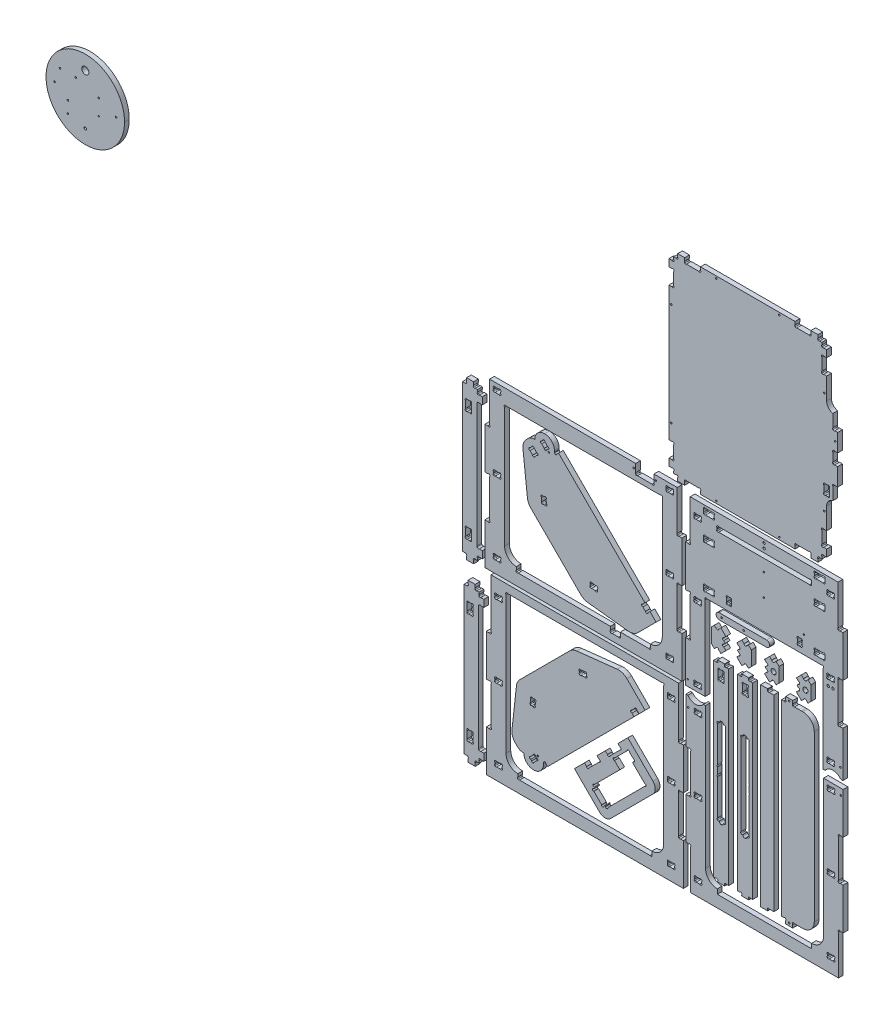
SolidWorks part; units mm, degrees
ref_plane "Plan de face" through (0, 0, 0) normal (0, 0, 1) x (1, 0, 0)
ref_plane "Plan de dessus" through (0, 0, 0) normal (0, 1, 0) x (1, 0, 0)
ref_plane "Plan de droite" through (0, 0, 0) normal (1, 0, 0) x (0, 0, -1)
sketch "Model" plane through (0, 0, 0) normal (0, 0, 1) x (1, 0, 0)
  line L0 (2110.7773, 190.5964) -> (2109.7418, 190.5964)
  line L1 (2102.6707, 187.6675) -> (2100.0908, 185.0876)
  line L2 (2095.7892, 172.8245) -> (2101.483, 121.5797)
  line L3 (2105.7847, 112.6296) -> (2169.0542, 49.3601)
  line L4 (2178.0043, 45.0585) -> (2229.2491, 39.3646)
  line L5 (2241.5122, 43.6662) -> (2264.6987, 66.8527)
  line L6 (2264.6987, 66.8527) -> (2256.9205, 74.6309)
  line L7 (2256.9205, 74.6309) -> (2254.2278, 71.9383)
  line L8 (2251.1278, 71.9383) -> (2247.8639, 75.2022)
  line L9 (2247.8639, 78.3022) -> (2250.5565, 80.9949)
  line L10 (2250.5565, 80.9949) -> (2140.955, 190.5964)
  line L11 (2140.955, 190.5964) -> (2138.9694, 188.6109)
  line L12 (2135.8694, 188.6109) -> (2135.6517, 188.8286)
  line L13 (2119.6514, 126.5979) -> (2119.1416, 131.1856)
  line L14 (2121.0782, 133.6063) -> (2122.6842, 133.7847)
  line L15 (2125.1049, 131.8482) -> (2125.6147, 127.2605)
  line L16 (2123.6781, 124.8398) -> (2122.0721, 124.6613)
  line L17 (2183.6851, 69.1901) -> (2188.2728, 68.6803)
  line L18 (2190.2093, 66.2596) -> (2190.0309, 64.6536)
  line L19 (2187.6102, 62.717) -> (2183.0225, 63.2268)
  line L20 (2181.0859, 65.6475) -> (2181.2644, 67.2535)
  line L21 (2123.7666, 194.3497) -> (2127.0306, 191.0857)
  line L22 (2127.0306, 187.9857) -> (2125.888, 186.8431)
  line L23 (2122.788, 186.8431) -> (2119.524, 190.1071)
  line L24 (2119.524, 193.2071) -> (2120.6666, 194.3497)
  line L25 (2109.984, 180.5671) -> (2113.248, 177.3031)
  line L26 (2113.248, 174.2031) -> (2111.1075, 172.0627)
  line L27 (2108.0075, 172.0627) -> (2104.7436, 175.3266)
  line L28 (2104.7436, 178.4266) -> (2106.884, 180.5671)
  line L29 (2259.9927, 67.3161) -> (2234.4782, 41.782)
  line L30 (2234.4782, 41.782) -> (2174.0683, 48.4587)
  line L31 (2174.0683, 48.4587) -> (2104.95, 117.7599)
  line L32 (2104.95, 117.7599) -> (2098.1492, 178.8558)
  line L33 (2098.1492, 178.8558) -> (2106.6943, 187.4008)
  line L34 (2106.6943, 187.4008) -> (2121.156, 188.4751)
  line L35 (2192.3959, -119.9378) -> (2189.7032, -117.2451)
  line L36 (2189.7032, -117.2451) -> (2200.3098, -106.6385)
  line L37 (2200.3098, -106.6385) -> (2203.0025, -109.3312)
  line L38 (2206.1025, -109.3312) -> (2218.9124, -96.5213)
  line L39 (2218.9124, -93.4213) -> (2216.2198, -90.7286)
  line L40 (2216.2198, -90.7286) -> (2228.8453, -78.0215)
  line L41 (2228.8453, -78.0215) -> (2260.6651, -109.8413)
  line L42 (2260.6651, -123.9834) -> (2207.0803, -177.6498)
  line L43 (2192.9382, -177.6498) -> (2161.1184, -145.83)
  line L44 (2161.1184, -145.83) -> (2173.7933, -133.155)
  line L45 (2173.7933, -133.155) -> (2176.486, -135.8477)
  line L46 (2179.586, -135.8477) -> (2192.3959, -123.0378)
  line L47 (2051.2882, 70.6746) -> (2047.4802, 70.6746)
  line L48 (2047.4802, 70.6746) -> (2047.4802, 18.1746)
  line L49 (2047.4802, 18.1746) -> (2072.4802, 18.1746)
  line L50 (2072.4802, 18.1746) -> (2272.4825, 18.1746)
  line L51 (2272.4825, 18.1746) -> (2297.4825, 18.1746)
  line L52 (2297.4825, 18.1746) -> (2297.4825, 70.6746)
  line L53 (2297.4825, 70.6746) -> (2293.6746, 70.6746)
  line L54 (2291.4825, 72.8666) -> (2291.4825, 120.9826)
  line L55 (2293.6746, 123.1746) -> (2297.4825, 123.1746)
  line L56 (2297.4825, 123.1746) -> (2297.4825, 175.6746)
  line L57 (2297.4825, 175.6746) -> (2293.6746, 175.6746)
  line L58 (2291.4825, 177.8666) -> (2291.4825, 218.1746)
  line L59 (2291.4825, 218.1746) -> (2291.4825, 228.1746)
  line L60 (2291.4825, 228.1746) -> (2261.9085, 228.1746)
  line L61 (2261.9085, 228.1746) -> (2261.9085, 218.0683)
  line L62 (2259.7164, 215.8762) -> (2241.0005, 215.8762)
  line L63 (2238.8084, 218.0683) -> (2238.8084, 228.1746)
  line L64 (2238.8084, 228.1746) -> (2053.4802, 228.1746)
  line L65 (2053.4802, 228.1746) -> (2053.4802, 218.1746)
  line L66 (2053.4802, 218.1746) -> (2053.4802, 177.8666)
  line L67 (2051.2882, 175.6746) -> (2047.4802, 175.6746)
  line L68 (2047.4802, 175.6746) -> (2047.4802, 123.1746)
  line L69 (2047.4802, 123.1746) -> (2051.2882, 123.1746)
  line L70 (2053.4802, 120.9826) -> (2053.4802, 72.8666)
  line L71 (2397.177, 64.4112) -> (2397.177, -179.5888)
  line L72 (2397.177, -179.5888) -> (2406.177, -179.5888)
  line L73 (2406.177, -179.5888) -> (2406.177, -178.7102)
  line L74 (2408.2983, -176.5889) -> (2413.9379, -176.5889)
  line L75 (2413.9379, -176.5889) -> (2413.9379, 61.4113)
  line L76 (2413.9379, 61.4113) -> (2408.2983, 61.4113)
  line L77 (2406.177, 63.5324) -> (2406.177, 64.4112)
  line L78 (2406.177, 64.4112) -> (2397.177, 64.4112)
  line L79 (2426.8343, 61.4113) -> (2423.9557, 61.4113)
  line L80 (2423.9557, 61.4113) -> (2423.9557, -176.5889)
  line L81 (2423.9557, -176.5889) -> (2426.8343, -176.5889)
  line L82 (2428.9557, -178.7102) -> (2428.9557, -182.5888)
  line L83 (2428.9557, -182.5888) -> (2437.9557, -182.5888)
  line L84 (2437.9557, -182.5888) -> (2437.9557, -178.7102)
  line L85 (2440.077, -176.5889) -> (2444.7718, -176.5889)
  line L86 (2444.7718, -176.5889) -> (2445.7718, -176.5889)
  line L87 (2445.7718, -176.5889) -> (2448.9557, -176.5889)
  line L88 (2448.9557, -176.5889) -> (2450.713, -176.5889)
  line L89 (2465.2718, -162.03) -> (2465.2718, 46.8524)
  line L90 (2450.713, 61.4113) -> (2448.9557, 61.4113)
  line L91 (2448.9557, 61.4113) -> (2445.7718, 61.4113)
  line L92 (2445.7718, 61.4113) -> (2444.7718, 61.4113)
  line L93 (2444.7718, 61.4113) -> (2440.077, 61.4113)
  line L94 (2437.9557, 63.5324) -> (2437.9557, 67.4112)
  line L95 (2437.9557, 67.4112) -> (2428.9557, 67.4112)
  line L96 (2428.9557, 67.4112) -> (2428.9557, 63.5324)
  line L97 (2096.8563, -160.6956) -> (2095.8208, -160.6956)
  line L98 (2088.7497, -157.7667) -> (2086.1699, -155.1868)
  line L99 (2081.8682, -142.9237) -> (2087.5621, -91.6789)
  line L100 (2091.8637, -82.7288) -> (2155.1332, -19.4593)
  line L101 (2164.0834, -15.1576) -> (2215.3282, -9.4638)
  line L102 (2227.5912, -13.7654) -> (2250.7777, -36.9519)
  line L103 (2250.7777, -36.9519) -> (2242.9995, -44.7301)
  line L104 (2242.9995, -44.7301) -> (2240.3069, -42.0374)
  line L105 (2237.2069, -42.0374) -> (2233.9429, -45.3014)
  line L106 (2233.9429, -48.4014) -> (2236.6356, -51.094)
  line L107 (2236.6356, -51.094) -> (2127.034, -160.6956)
  line L108 (2127.034, -160.6956) -> (2125.0485, -158.7101)
  line L109 (2121.9485, -158.7101) -> (2121.7307, -158.9278)
  line L110 (2105.7304, -96.6971) -> (2105.2207, -101.2848)
  line L111 (2107.1572, -103.7055) -> (2108.7633, -103.8839)
  line L112 (2111.184, -101.9474) -> (2111.6937, -97.3597)
  line L113 (2109.7571, -94.939) -> (2108.1511, -94.7605)
  line L114 (2169.7641, -39.2893) -> (2174.3518, -38.7795)
  line L115 (2176.2884, -36.3588) -> (2176.1099, -34.7528)
  line L116 (2173.6892, -32.8162) -> (2169.1015, -33.326)
  line L117 (2167.165, -35.7467) -> (2167.3434, -37.3527)
  line L118 (2109.8457, -164.4489) -> (2113.1096, -161.1849)
  line L119 (2113.1096, -158.0849) -> (2111.967, -156.9423)
  line L120 (2108.867, -156.9423) -> (2105.603, -160.2063)
  line L121 (2105.603, -163.3063) -> (2106.7457, -164.4489)
  line L122 (2246.0717, -37.4153) -> (2220.5573, -11.8812)
  line L123 (2220.5573, -11.8812) -> (2160.1473, -18.5579)
  line L124 (2160.1473, -18.5579) -> (2091.029, -87.8591)
  line L125 (2091.029, -87.8591) -> (2084.2282, -148.955)
  line L126 (2084.2282, -148.955) -> (2092.7733, -157.5)
  line L127 (2092.7733, -157.5) -> (2107.235, -158.5743)
  line L128 (2024.9826, -172.2811) -> (2024.9826, -181.1304)
  line L129 (2027.1746, -183.3224) -> (2030.2017, -183.3224)
  line L130 (2032.3937, -181.1304) -> (2032.3937, -172.2811)
  line L131 (2030.2017, -170.0891) -> (2027.1746, -170.0891)
  line L132 (2024.9826, -31.9928) -> (2024.9826, -40.842)
  line L133 (2027.1746, -43.0341) -> (2030.2017, -43.0341)
  line L134 (2032.3937, -40.842) -> (2032.3937, -31.9928)
  line L135 (2030.2017, -29.8007) -> (2027.1746, -29.8007)
  line L136 (2021.1891, -194.352) -> (2021.1887, -199.552)
  line L137 (2021.1887, -199.552) -> (2024.6416, -199.5522)
  line L138 (2026.1886, -202.5443) -> (2026.1883, -206.3523)
  line L139 (2026.1883, -206.3523) -> (2035.1884, -206.3528)
  line L140 (2035.1884, -206.3528) -> (2035.1885, -202.5448)
  line L141 (2037.3807, -200.3529) -> (2040.1887, -200.3531)
  line L142 (2040.1887, -200.3531) -> (2040.1888, -197.5451)
  line L143 (2042.381, -195.3532) -> (2046.189, -195.3534)
  line L144 (2046.189, -195.3534) -> (2046.1895, -186.3534)
  line L145 (2046.1895, -186.3534) -> (2042.3816, -186.3532)
  line L146 (2039.3896, -184.8059) -> (2039.3896, -184.3053)
  line L147 (2039.3896, -184.3053) -> (2039.3965, -184.302)
  line L148 (2039.3965, -184.302) -> (2039.3965, -27.8103)
  line L149 (2042.3816, -26.3519) -> (2046.1895, -26.3516)
  line L150 (2046.1895, -26.3516) -> (2046.189, -17.3516)
  line L151 (2046.189, -17.3516) -> (2042.381, -17.3519)
  line L152 (2040.1888, -15.16) -> (2040.1887, -12.352)
  line L153 (2040.1887, -12.352) -> (2037.3807, -12.3521)
  line L154 (2035.1885, -10.1602) -> (2035.1884, -6.3523)
  line L155 (2035.1884, -6.3523) -> (2026.1883, -6.3528)
  line L156 (2026.1883, -6.3528) -> (2026.1886, -10.1608)
  line L157 (2024.6416, -13.1529) -> (2021.1887, -13.1531)
  line L158 (2021.1887, -13.1531) -> (2021.1891, -18.3531)
  line L159 (2021.1891, -18.3531) -> (2021.1891, -194.352)
  line L160 (2349.6678, -61.8906) -> (2349.6678, -53.287)
  line L161 (2347.4758, -51.095) -> (2344.5279, -51.095)
  line L162 (2342.3359, -53.287) -> (2342.3359, -61.8906)
  line L163 (2344.5279, -64.0826) -> (2347.4758, -64.0826)
  line L164 (2494.9366, 330.2781) -> (2491.1286, 330.2781)
  line L165 (2488.9366, 328.0861) -> (2488.9366, 312.3492)
  line L166 (2480.9366, 302.5512) -> (2480.9366, 275.2781)
  line L167 (2480.9366, 275.2781) -> (2477.1286, 275.2781)
  line L168 (2474.9366, 273.0861) -> (2474.9366, 257.4701)
  line L169 (2477.1286, 255.2781) -> (2480.9366, 255.2781)
  line L170 (2480.9366, 255.2781) -> (2480.9366, 246.2781)
  line L171 (2480.9366, 246.2781) -> (2477.1286, 246.2781)
  line L172 (2474.9366, 244.0861) -> (2474.9366, 241.2781)
  line L173 (2474.9366, 241.2781) -> (2472.1286, 241.2781)
  line L174 (2469.9366, 239.0861) -> (2469.9366, 235.2781)
  line L175 (2469.9366, 235.2781) -> (2460.9366, 235.2781)
  line L176 (2460.9366, 235.2781) -> (2460.9366, 239.0861)
  line L177 (2458.7445, 241.2781) -> (2443.1286, 241.2781)
  line L178 (2440.9366, 239.0861) -> (2440.9366, 235.2781)
  line L179 (2440.9366, 235.2781) -> (2320.9366, 235.2781)
  line L180 (2320.9366, 235.2781) -> (2320.9366, 239.0861)
  line L181 (2318.7445, 241.2781) -> (2303.1286, 241.2781)
  line L182 (2300.9366, 239.0861) -> (2300.9366, 235.2781)
  line L183 (2300.9366, 235.2781) -> (2291.9366, 235.2781)
  line L184 (2291.9366, 235.2781) -> (2291.9366, 239.0861)
  line L185 (2289.7445, 241.2781) -> (2286.9366, 241.2781)
  line L186 (2286.9366, 241.2781) -> (2286.9366, 244.0861)
  line L187 (2284.7445, 246.2781) -> (2280.9366, 246.2781)
  line L188 (2280.9366, 246.2781) -> (2280.9366, 255.2781)
  line L189 (2280.9366, 255.2781) -> (2284.7445, 255.2781)
  line L190 (2286.9366, 257.4701) -> (2286.9366, 273.0861)
  line L191 (2284.7445, 275.2781) -> (2280.9366, 275.2781)
  line L192 (2280.9366, 275.2781) -> (2280.9366, 445.2781)
  line L193 (2280.9366, 445.2781) -> (2284.7445, 445.2781)
  line L194 (2286.9366, 447.4701) -> (2286.9366, 463.0861)
  line L195 (2284.7445, 465.2781) -> (2280.9366, 465.2781)
  line L196 (2280.9366, 465.2781) -> (2280.9366, 474.2781)
  line L197 (2280.9366, 474.2781) -> (2284.7445, 474.2781)
  line L198 (2286.9366, 476.4701) -> (2286.9366, 479.2781)
  line L199 (2286.9366, 479.2781) -> (2289.7445, 479.2781)
  line L200 (2291.9366, 481.4701) -> (2291.9366, 485.2781)
  line L201 (2291.9366, 485.2781) -> (2300.9366, 485.2781)
  line L202 (2300.9366, 485.2781) -> (2300.9366, 481.4701)
  line L203 (2303.1286, 479.2781) -> (2318.7445, 479.2781)
  line L204 (2320.9366, 481.4701) -> (2320.9366, 485.2781)
  line L205 (2320.9366, 485.2781) -> (2440.9366, 485.2781)
  line L206 (2440.9366, 485.2781) -> (2440.9366, 481.4701)
  line L207 (2443.1286, 479.2781) -> (2458.7445, 479.2781)
  line L208 (2460.9366, 481.4701) -> (2460.9366, 485.2781)
  line L209 (2460.9366, 485.2781) -> (2469.9366, 485.2781)
  line L210 (2469.9366, 485.2781) -> (2469.9366, 481.4701)
  line L211 (2472.1286, 479.2781) -> (2474.9366, 479.2781)
  line L212 (2474.9366, 479.2781) -> (2474.9366, 476.4701)
  line L213 (2477.1286, 474.2781) -> (2480.9366, 474.2781)
  line L214 (2480.9366, 474.2781) -> (2480.9366, 465.2781)
  line L215 (2480.9366, 465.2781) -> (2477.1286, 465.2781)
  line L216 (2474.9366, 463.0861) -> (2474.9366, 447.4701)
  line L217 (2477.1286, 445.2781) -> (2480.9366, 445.2781)
  line L218 (2480.9366, 445.2781) -> (2480.9366, 418.005)
  line L219 (2488.9366, 408.207) -> (2488.9366, 392.4701)
  line L220 (2491.1286, 390.2781) -> (2494.9366, 390.2781)
  line L221 (2494.9366, 390.2781) -> (2494.9366, 367.7781)
  line L222 (2494.9366, 367.7781) -> (2491.1286, 367.7781)
  line L223 (2488.9366, 365.5861) -> (2488.9366, 354.9701)
  line L224 (2491.1286, 352.7781) -> (2494.9366, 352.7781)
  line L225 (2494.9366, 352.7781) -> (2494.9366, 330.2781)
  line L226 (2286.9366, 479.2525) -> (2474.9366, 479.2525)
  line L227 (2474.9366, 479.2525) -> (2474.9366, 241.2781)
  line L228 (2474.9366, 241.2781) -> (2286.9366, 241.2781)
  line L229 (2286.9366, 241.2781) -> (2286.9366, 479.2525)
  line L230 (2477.3874, 323.7689) -> (2477.3874, 315.6252)
  line L231 (2479.5795, 313.4332) -> (2482.2537, 313.4332)
  line L232 (2484.4458, 315.6252) -> (2484.4458, 323.7689)
  line L233 (2482.2537, 325.961) -> (2479.5795, 325.961)
  line L234 (2067.1066, -187.2653) -> (2062.4907, -187.2653)
  line L235 (2060.2987, -189.4573) -> (2060.2987, -191.0732)
  line L236 (2062.4907, -193.2653) -> (2067.1066, -193.2653)
  line L237 (2069.2987, -191.0732) -> (2069.2987, -189.4573)
  line L238 (2281.4907, -187.2653) -> (2286.1066, -187.2653)
  line L239 (2288.2987, -189.4573) -> (2288.2987, -191.0732)
  line L240 (2286.1066, -193.2653) -> (2281.4907, -193.2653)
  line L241 (2279.2987, -191.0732) -> (2279.2987, -189.4573)
  line L242 (2484.1661, -187.2762) -> (2488.782, -187.2762)
  line L243 (2490.974, -189.4682) -> (2490.974, -191.0841)
  line L244 (2488.782, -193.2762) -> (2484.1661, -193.2762)
  line L245 (2481.974, -191.0841) -> (2481.974, -189.4682)
  line L246 (2484.1661, -3.3762) -> (2488.782, -3.3762)
  line L247 (2490.974, -5.5682) -> (2490.974, -7.1841)
  line L248 (2488.782, -9.3762) -> (2484.1661, -9.3762)
  line L249 (2481.974, -7.1841) -> (2481.974, -5.5682)
  line L250 (2342.3323, -193.2762) -> (2342.3323, -187.2762)
  line L251 (2327.3323, -172.2762) -> (2327.3323, 6.6238)
  line L252 (2327.3323, 6.6238) -> (2324.8323, 6.6238)
  line L253 (2304.8323, 6.6238) -> (2302.3323, 6.6238)
  line L254 (2302.3323, 6.6238) -> (2302.3323, -50.8762)
  line L255 (2302.3323, -50.8762) -> (2306.1403, -50.8762)
  line L256 (2308.3323, -53.0682) -> (2308.3323, -101.1841)
  line L257 (2306.1403, -103.3762) -> (2302.3323, -103.3762)
  line L258 (2302.3323, -103.3762) -> (2302.3323, -155.8762)
  line L259 (2302.3323, -155.8762) -> (2306.1403, -155.8762)
  line L260 (2308.3323, -158.0682) -> (2308.3323, -208.3762)
  line L261 (2308.3323, -208.3762) -> (2327.3323, -208.3762)
  line L262 (2327.3323, -208.3762) -> (2476.974, -208.3762)
  line L263 (2476.974, -208.3762) -> (2495.974, -208.3762)
  line L264 (2495.974, -208.3762) -> (2495.974, -158.0682)
  line L265 (2498.1661, -155.8762) -> (2501.974, -155.8762)
  line L266 (2501.974, -155.8762) -> (2501.974, -103.3762)
  line L267 (2501.974, -103.3762) -> (2498.1661, -103.3762)
  line L268 (2495.974, -101.1841) -> (2495.974, -53.0682)
  line L269 (2498.1661, -50.8762) -> (2501.974, -50.8762)
  line L270 (2501.974, -50.8762) -> (2501.974, 1.6238)
  line L271 (2501.974, 1.6238) -> (2476.974, 1.6238)
  line L272 (2476.974, 1.6238) -> (2476.974, -172.2762)
  line L273 (2461.974, -187.2762) -> (2461.974, -193.2762)
  line L274 (2461.974, -193.2762) -> (2342.3323, -193.2762)
  line L275 (2320.1403, -187.2762) -> (2315.5243, -187.2762)
  line L276 (2313.3323, -189.4682) -> (2313.3323, -191.0841)
  line L277 (2315.5243, -193.2762) -> (2320.1403, -193.2762)
  line L278 (2322.3323, -191.0841) -> (2322.3323, -189.4682)
  line L279 (2320.1403, -3.3762) -> (2315.5243, -3.3762)
  line L280 (2313.3323, -5.5682) -> (2313.3323, -7.1841)
  line L281 (2315.5243, -9.3762) -> (2320.1403, -9.3762)
  line L282 (2322.3323, -7.1841) -> (2322.3323, -5.5682)
  line L283 (2279.6745, 39.2746) -> (2284.2905, 39.2746)
  line L284 (2286.4825, 37.0826) -> (2286.4825, 35.4666)
  line L285 (2284.2905, 33.2746) -> (2279.6745, 33.2746)
  line L286 (2277.4825, 35.4666) -> (2277.4825, 37.0826)
  line L287 (2279.6745, 223.1746) -> (2284.2905, 223.1746)
  line L288 (2286.4825, 220.9826) -> (2286.4825, 219.3666)
  line L289 (2284.2905, 217.1746) -> (2279.6745, 217.1746)
  line L290 (2277.4825, 219.3666) -> (2277.4825, 220.9826)
  line L291 (2065.2882, 39.2746) -> (2060.6722, 39.2746)
  line L292 (2058.4802, 37.0826) -> (2058.4802, 35.4666)
  line L293 (2060.6722, 33.2746) -> (2065.2882, 33.2746)
  line L294 (2067.4802, 35.4666) -> (2067.4802, 37.0826)
  line L295 (2065.2882, 223.1746) -> (2060.6722, 223.1746)
  line L296 (2058.4802, 220.9826) -> (2058.4802, 219.3666)
  line L297 (2060.6722, 217.1746) -> (2065.2882, 217.1746)
  line L298 (2067.4802, 219.3666) -> (2067.4802, 220.9826)
  line L299 (2295.4907, -103.3653) -> (2299.2987, -103.3653)
  line L300 (2299.2987, -103.3653) -> (2299.2987, -50.8653)
  line L301 (2299.2987, -50.8653) -> (2295.4907, -50.8653)
  line L302 (2293.2987, -48.6732) -> (2293.2987, 4.1347)
  line L303 (2293.2987, 4.1347) -> (2293.2987, 14.1347)
  line L304 (2293.2987, 14.1347) -> (2274.2987, 14.1347)
  line L305 (2274.2987, 14.1347) -> (2074.2987, 14.1347)
  line L306 (2074.2987, 14.1347) -> (2055.2987, 14.1347)
  line L307 (2055.2987, 14.1347) -> (2055.2987, 4.1347)
  line L308 (2055.2987, 4.1347) -> (2055.2987, -48.6732)
  line L309 (2053.1066, -50.8653) -> (2049.2987, -50.8653)
  line L310 (2049.2987, -50.8653) -> (2049.2987, -103.3653)
  line L311 (2049.2987, -103.3653) -> (2053.1066, -103.3653)
  line L312 (2055.2987, -105.5573) -> (2055.2987, -153.6732)
  line L313 (2053.1066, -155.8653) -> (2049.2987, -155.8653)
  line L314 (2049.2987, -155.8653) -> (2049.2987, -208.3653)
  line L315 (2049.2987, -208.3653) -> (2074.2987, -208.3653)
  line L316 (2074.2987, -208.3653) -> (2274.2987, -208.3653)
  line L317 (2274.2987, -208.3653) -> (2299.2987, -208.3653)
  line L318 (2299.2987, -208.3653) -> (2299.2987, -155.8653)
  line L319 (2299.2987, -155.8653) -> (2295.4907, -155.8653)
  line L320 (2293.2987, -153.6732) -> (2293.2987, -105.5573)
  line L321 (2274.2987, 4.1255) -> (2274.2874, 4.1347)
  line L322 (2272.1066, 4.1347) -> (2272.0527, 4.1347)
  line L323 (2272.0527, 4.1347) -> (2076.5446, 4.1347)
  line L324 (2076.5446, 4.1347) -> (2076.4907, 4.1347)
  line L325 (2074.31, 4.1347) -> (2074.2987, 4.1255)
  line L326 (2074.2987, 1.9335) -> (2074.2987, -172.2653)
  line L327 (2089.2987, -187.2653) -> (2089.2987, -191.0732)
  line L328 (2091.4907, -193.2653) -> (2257.1066, -193.2653)
  line L329 (2259.2987, -191.0732) -> (2259.2987, -187.2653)
  line L330 (2274.2987, -172.2653) -> (2274.2987, 1.9335)
  line L331 (2385.431, 96.7088) -> (2385.4321, 78.324)
  line L332 (2385.4321, 78.324) -> (2381.7553, 74.6469)
  line L333 (2381.7553, 74.6469) -> (2379.3137, 77.0883)
  line L334 (2376.104, 76.0664) -> (2373.4116, 73.3736)
  line L335 (2373.4116, 73.3736) -> (2367.0472, 79.7372)
  line L336 (2367.0472, 79.7372) -> (2369.7397, 82.43)
  line L337 (2369.7395, 85.53) -> (2367.7539, 87.5154)
  line L338 (2367.7539, 87.5154) -> (2369.7393, 89.501)
  line L339 (2369.7391, 92.601) -> (2367.0463, 95.2935)
  line L340 (2367.0463, 95.2935) -> (2373.4099, 101.6579)
  line L341 (2373.4099, 101.6579) -> (2376.1027, 98.9654)
  line L342 (2379.3125, 97.9439) -> (2381.7539, 100.3855)
  line L343 (2381.7539, 100.3855) -> (2385.431, 96.7088)
  line L344 (2334.8114, 78.3226) -> (2334.8103, 96.7074)
  line L345 (2334.8103, 96.7074) -> (2338.487, 100.3846)
  line L346 (2338.487, 100.3846) -> (2340.9287, 97.9432)
  line L347 (2344.1383, 98.9651) -> (2346.8308, 101.6579)
  line L348 (2346.8308, 101.6579) -> (2353.1952, 95.2943)
  line L349 (2353.1952, 95.2943) -> (2350.5027, 92.6015)
  line L350 (2350.5028, 89.5015) -> (2352.4885, 87.516)
  line L351 (2352.4885, 87.516) -> (2350.5031, 85.5304)
  line L352 (2350.5033, 82.4304) -> (2353.196, 79.7379)
  line L353 (2353.196, 79.7379) -> (2346.8325, 73.3736)
  line L354 (2346.8325, 73.3736) -> (2344.1397, 76.0661)
  line L355 (2340.9299, 77.0876) -> (2338.4885, 74.6459)
  line L356 (2338.4885, 74.6459) -> (2334.8114, 78.3226)
  line L357 (2420.5659, 96.1295) -> (2420.567, 77.7447)
  line L358 (2420.567, 77.7447) -> (2416.8902, 74.0676)
  line L359 (2416.8902, 74.0676) -> (2414.4485, 76.509)
  line L360 (2411.2389, 75.4871) -> (2408.5464, 72.7943)
  line L361 (2408.5464, 72.7943) -> (2402.1821, 79.1579)
  line L362 (2402.1821, 79.1579) -> (2404.8746, 81.8507)
  line L363 (2404.8744, 84.9507) -> (2402.8888, 86.9361)
  line L364 (2402.8888, 86.9361) -> (2404.8742, 88.9217)
  line L365 (2404.874, 92.0217) -> (2402.1812, 94.7142)
  line L366 (2402.1812, 94.7142) -> (2408.5448, 101.0786)
  line L367 (2408.5448, 101.0786) -> (2411.2376, 98.3861)
  line L368 (2414.4473, 97.3646) -> (2416.8887, 99.8062)
  line L369 (2416.8887, 99.8062) -> (2420.5659, 96.1295)
  line L370 (2185.7384, -158.4095) -> (2195.5758, -168.2469)
  line L371 (2198.4737, -168.2252) -> (2199.8836, -166.8153)
  line L372 (2199.8836, -166.8153) -> (2200.5434, -167.4752)
  line L373 (2203.4217, -167.5199) -> (2250.2962, -120.6454)
  line L374 (2250.311, -117.7487) -> (2234.7814, -102.219)
  line L375 (2234.7814, -102.219) -> (2236.0377, -100.9628)
  line L376 (2236.0377, -97.8627) -> (2231.0088, -92.8338)
  line L377 (2227.9087, -92.8338) -> (2212.0779, -108.6592)
  line L378 (2211.9646, -111.5757) -> (2218.6947, -118.3057)
  line L379 (2218.6947, -118.3057) -> (2186.4436, -150.5568)
  line L380 (2186.5101, -153.4419) -> (2187.1556, -154.0874)
  line L381 (2187.1556, -154.0874) -> (2185.7382, -155.5048)
  line L382 (2067.1066, -95.3153) -> (2062.4907, -95.3153)
  line L383 (2060.2987, -97.5073) -> (2060.2987, -99.1232)
  line L384 (2062.4907, -101.3153) -> (2067.1066, -101.3153)
  line L385 (2069.2987, -99.1232) -> (2069.2987, -97.5073)
  line L386 (2281.4907, -95.3153) -> (2286.1066, -95.3153)
  line L387 (2288.2987, -97.5073) -> (2288.2987, -99.1232)
  line L388 (2286.1066, -101.3153) -> (2281.4907, -101.3153)
  line L389 (2279.2987, -99.1232) -> (2279.2987, -97.5073)
  line L390 (2279.6745, 125.2246) -> (2284.2905, 125.2246)
  line L391 (2286.4825, 127.4166) -> (2286.4825, 129.0326)
  line L392 (2284.2905, 131.2246) -> (2279.6745, 131.2246)
  line L393 (2277.4825, 129.0326) -> (2277.4825, 127.4166)
  line L394 (2488.7713, -95.3257) -> (2484.1554, -95.3257)
  line L395 (2481.9633, -97.5177) -> (2481.9633, -99.1337)
  line L396 (2484.1554, -101.3257) -> (2488.7713, -101.3257)
  line L397 (2490.9633, -99.1337) -> (2490.9633, -97.5177)
  line L398 (2320.1291, -95.3257) -> (2315.5132, -95.3257)
  line L399 (2313.3211, -97.5177) -> (2313.3211, -99.1337)
  line L400 (2315.5132, -101.3257) -> (2320.1291, -101.3257)
  line L401 (2322.3211, -99.1337) -> (2322.3211, -97.5177)
  line L402 (2065.2905, 125.2246) -> (2060.6745, 125.2246)
  line L403 (2058.4825, 127.4166) -> (2058.4825, 129.0326)
  line L404 (2060.6745, 131.2246) -> (2065.2905, 131.2246)
  line L405 (2067.4825, 129.0326) -> (2067.4825, 127.4166)
  line L406 (2074.7285, 209.0719) -> (2074.6746, 209.0719)
  line L407 (2072.4938, 209.0719) -> (2072.4825, 209.0627)
  line L408 (2072.4825, 206.8707) -> (2072.4825, 54.2746)
  line L409 (2087.4826, 39.2746) -> (2087.4826, 35.4666)
  line L410 (2089.6745, 33.2746) -> (2206.7997, 33.2746)
  line L411 (2206.7997, 33.2746) -> (2206.7997, 28.7967)
  line L412 (2208.9916, 26.6046) -> (2217.1354, 26.6046)
  line L413 (2219.3274, 28.7967) -> (2219.3274, 33.2746)
  line L414 (2219.3274, 33.2746) -> (2255.2905, 33.2746)
  line L415 (2257.4825, 35.4666) -> (2257.4825, 39.2746)
  line L416 (2272.4825, 54.2746) -> (2272.4825, 206.8707)
  line L417 (2272.4825, 209.0627) -> (2272.4712, 209.0719)
  line L418 (2270.2905, 209.0719) -> (2270.2365, 209.0719)
  line L419 (2270.2365, 209.0719) -> (2231.3896, 209.0719)
  line L420 (2404.6925, 109.2838) -> (2344.8091, 109.2838)
  line L421 (2344.8091, 117.2838) -> (2404.6925, 117.2838)
  line L422 (2022.9838, 49.1999) -> (2022.9838, 40.3507)
  line L423 (2025.1758, 38.1586) -> (2028.2028, 38.1586)
  line L424 (2030.3949, 40.3507) -> (2030.3949, 49.1999)
  line L425 (2028.2028, 51.392) -> (2025.1758, 51.392)
  line L426 (2022.9838, 189.4883) -> (2022.9838, 180.6391)
  line L427 (2025.1758, 178.447) -> (2028.2028, 178.447)
  line L428 (2030.3949, 180.6391) -> (2030.3949, 189.4883)
  line L429 (2028.2028, 191.6804) -> (2025.1758, 191.6804)
  line L430 (2019.1902, 27.1291) -> (2019.1899, 21.9291)
  line L431 (2019.1899, 21.9291) -> (2022.6427, 21.9289)
  line L432 (2024.1897, 18.9368) -> (2024.1895, 15.1288)
  line L433 (2024.1895, 15.1288) -> (2033.1895, 15.1283)
  line L434 (2033.1895, 15.1283) -> (2033.1897, 18.9363)
  line L435 (2035.3818, 21.1282) -> (2038.1898, 21.128)
  line L436 (2038.1898, 21.128) -> (2038.19, 23.936)
  line L437 (2040.3822, 26.1279) -> (2044.1901, 26.1277)
  line L438 (2044.1901, 26.1277) -> (2044.1907, 35.1277)
  line L439 (2044.1907, 35.1277) -> (2040.3827, 35.1279)
  line L440 (2037.3907, 36.6752) -> (2037.3907, 37.1758)
  line L441 (2037.3907, 37.1758) -> (2037.3976, 37.1791)
  line L442 (2037.3976, 37.1791) -> (2037.3976, 193.6708)
  line L443 (2040.3827, 195.1292) -> (2044.1907, 195.1295)
  line L444 (2044.1907, 195.1295) -> (2044.1901, 204.1294)
  line L445 (2044.1901, 204.1294) -> (2040.3822, 204.1292)
  line L446 (2038.19, 206.3211) -> (2038.1898, 209.1291)
  line L447 (2038.1898, 209.1291) -> (2035.3818, 209.1289)
  line L448 (2033.1897, 211.3208) -> (2033.1895, 215.1288)
  line L449 (2033.1895, 215.1288) -> (2024.1895, 215.1283)
  line L450 (2024.1895, 215.1283) -> (2024.1897, 211.3203)
  line L451 (2022.6427, 208.3282) -> (2019.1899, 208.328)
  line L452 (2019.1899, 208.328) -> (2019.1902, 203.128)
  line L453 (2019.1902, 203.128) -> (2019.1902, 27.1291)
  line L454 (2319.6704, 205.12) -> (2315.0545, 205.1203)
  line L455 (2312.8626, 207.3125) -> (2312.8627, 208.9284)
  line L456 (2315.0548, 211.1203) -> (2319.6708, 211.12)
  line L457 (2321.8627, 208.9279) -> (2321.8626, 207.3119)
  line L458 (2459.3321, 205.3179) -> (2344.032, 205.3182)
  line L459 (2341.8401, 207.5104) -> (2341.8402, 209.1263)
  line L460 (2344.0324, 211.3182) -> (2459.3325, 211.3179)
  line L461 (2461.5244, 209.1258) -> (2461.5243, 207.5098)
  line L462 (2319.6598, 21.22) -> (2315.0439, 21.2203)
  line L463 (2312.852, 23.4125) -> (2312.8521, 25.0284)
  line L464 (2315.0442, 27.2203) -> (2319.6602, 27.22)
  line L465 (2321.8521, 25.0279) -> (2321.852, 23.4119)
  line L466 (2483.6962, 205.1106) -> (2488.3122, 205.1103)
  line L467 (2490.5043, 207.3022) -> (2490.5044, 208.9182)
  line L468 (2488.3125, 211.1103) -> (2483.6966, 211.1106)
  line L469 (2481.5044, 208.9187) -> (2481.5043, 207.3027)
  line L470 (2483.6856, 21.2106) -> (2488.3016, 21.2103)
  line L471 (2490.4937, 23.4022) -> (2490.4938, 25.0182)
  line L472 (2488.3019, 27.2103) -> (2483.686, 27.2106)
  line L473 (2481.4938, 25.0187) -> (2481.4937, 23.4027)
  line L474 (2495.5054, 226.2099) -> (2476.5054, 226.211)
  line L475 (2476.5054, 226.211) -> (2326.8637, 226.2196)
  line L476 (2326.8637, 226.2196) -> (2307.8637, 226.2207)
  line L477 (2307.8637, 226.2207) -> (2307.8608, 175.9127)
  line L478 (2305.6686, 173.7208) -> (2301.8607, 173.7211)
  line L479 (2301.8607, 173.7211) -> (2301.8576, 121.2211)
  line L480 (2301.8576, 121.2211) -> (2305.6656, 121.2208)
  line L481 (2307.8575, 119.0287) -> (2307.8547, 70.9127)
  line L482 (2305.6626, 68.7208) -> (2301.8546, 68.7211)
  line L483 (2301.8546, 68.7211) -> (2301.8516, 16.2211)
  line L484 (2301.8516, 16.2211) -> (2326.8516, 16.2196)
  line L485 (2326.8516, 16.2196) -> (2326.8577, 122.4841)
  line L486 (2329.0502, 124.6756) -> (2474.3066, 124.6672)
  line L487 (2476.4994, 122.4762) -> (2476.493, 11.211)
  line L488 (2476.493, 11.211) -> (2478.993, 11.2109)
  line L489 (2498.993, 11.2097) -> (2501.493, 11.2096)
  line L490 (2501.493, 11.2096) -> (2501.4963, 68.7096)
  line L491 (2501.4963, 68.7096) -> (2497.6884, 68.7098)
  line L492 (2495.4965, 70.9019) -> (2495.4992, 119.0179)
  line L493 (2497.6914, 121.2098) -> (2501.4994, 121.2096)
  line L494 (2501.4994, 121.2096) -> (2501.5024, 173.7096)
  line L495 (2501.5024, 173.7096) -> (2497.6944, 173.7098)
  line L496 (2495.5025, 175.9019) -> (2495.5054, 226.2099)
  line L497 (2327.2844, 192.74) -> (2336.1337, 192.74)
  line L498 (2338.3257, 190.5479) -> (2338.3257, 187.5209)
  line L499 (2336.1337, 185.3289) -> (2327.2844, 185.3289)
  line L500 (2325.0924, 187.5209) -> (2325.0924, 190.5479)
  line L501 (2327.2844, 138.9102) -> (2336.1337, 138.9102)
  line L502 (2338.3257, 136.7182) -> (2338.3257, 133.6911)
  line L503 (2336.1337, 131.4991) -> (2327.2844, 131.4991)
  line L504 (2325.0924, 133.6911) -> (2325.0924, 136.7182)
  line L505 (2467.5728, 138.9102) -> (2476.4221, 138.9102)
  line L506 (2478.6141, 136.7182) -> (2478.6141, 133.6911)
  line L507 (2476.4221, 131.4991) -> (2467.5728, 131.4991)
  line L508 (2465.3808, 133.6911) -> (2465.3808, 136.7182)
  line L509 (2327.2844, 223.1751) -> (2336.1337, 223.1751)
  line L510 (2338.3257, 220.9831) -> (2338.3257, 217.9561)
  line L511 (2336.1337, 215.764) -> (2327.2844, 215.764)
  line L512 (2325.0924, 217.9561) -> (2325.0924, 220.9831)
  line L513 (2467.5728, 223.1751) -> (2476.4221, 223.1751)
  line L514 (2478.6141, 220.9831) -> (2478.6141, 217.9561)
  line L515 (2476.4221, 215.764) -> (2467.5728, 215.764)
  line L516 (2465.3808, 217.9561) -> (2465.3808, 220.9831)
  line L517 (2315.0547, 119.1704) -> (2319.6706, 119.1704)
  line L518 (2321.8626, 116.9783) -> (2321.8626, 115.3624)
  line L519 (2319.6706, 113.1704) -> (2315.0547, 113.1704)
  line L520 (2312.8626, 115.3624) -> (2312.8626, 116.9783)
  line L521 (2483.6969, 119.1704) -> (2488.3128, 119.1704)
  line L522 (2490.5048, 116.9783) -> (2490.5048, 115.3624)
  line L523 (2488.3128, 113.1704) -> (2483.6969, 113.1704)
  line L524 (2481.5048, 115.3624) -> (2481.5048, 116.9783)
  line L525 (2467.5534, 192.8479) -> (2476.4027, 192.8479)
  line L526 (2478.5947, 190.6558) -> (2478.5947, 187.6288)
  line L527 (2476.4027, 185.4367) -> (2467.5534, 185.4367)
  line L528 (2465.3614, 187.6288) -> (2465.3614, 190.6558)
  line L529 (2443.7039, 133.6911) -> (2443.7039, 138.3071)
  line L530 (2445.896, 140.4991) -> (2447.5119, 140.4991)
  line L531 (2449.7039, 138.3071) -> (2449.7039, 133.6911)
  line L532 (2447.5119, 131.4991) -> (2445.896, 131.4991)
  line L533 (2360.0025, 133.6911) -> (2360.0025, 138.3071)
  line L534 (2357.8105, 140.4991) -> (2356.1946, 140.4991)
  line L535 (2354.0025, 138.3071) -> (2354.0025, 133.6911)
  line L536 (2356.1946, 131.4991) -> (2357.8105, 131.4991)
  line L537 (2460.9885, 96.1295) -> (2460.9896, 77.7447)
  line L538 (2460.9896, 77.7447) -> (2457.3128, 74.0676)
  line L539 (2457.3128, 74.0676) -> (2454.8711, 76.509)
  line L540 (2451.6615, 75.4871) -> (2448.969, 72.7943)
  line L541 (2448.969, 72.7943) -> (2442.6047, 79.1579)
  line L542 (2442.6047, 79.1579) -> (2445.2972, 81.8507)
  line L543 (2445.297, 84.9507) -> (2443.3114, 86.9361)
  line L544 (2443.3114, 86.9361) -> (2445.2968, 88.9217)
  line L545 (2445.2966, 92.0217) -> (2442.6038, 94.7142)
  line L546 (2442.6038, 94.7142) -> (2448.9674, 101.0786)
  line L547 (2448.9674, 101.0786) -> (2451.6602, 98.3861)
  line L548 (2454.8699, 97.3646) -> (2457.3113, 99.8062)
  line L549 (2457.3113, 99.8062) -> (2460.9885, 96.1295)
  line L550 (2382.1353, -178.7808) -> (2382.1353, -179.5888)
  line L551 (2382.1353, -179.5888) -> (2373.1353, -179.5888)
  line L552 (2373.1353, -179.5888) -> (2373.1353, -178.7808)
  line L553 (2370.9433, -176.5888) -> (2368.1353, -176.5888)
  line L554 (2368.1353, -176.5888) -> (2368.1353, 61.4112)
  line L555 (2368.1353, 61.4112) -> (2370.9433, 61.4112)
  line L556 (2373.1353, 63.6032) -> (2373.1353, 64.4112)
  line L557 (2373.1353, 64.4112) -> (2382.1353, 64.4112)
  line L558 (2382.1353, 64.4112) -> (2382.1353, 63.6032)
  line L559 (2384.3274, 61.4112) -> (2387.1353, 61.4112)
  line L560 (2387.1353, 61.4112) -> (2387.1353, -176.5888)
  line L561 (2387.1353, -176.5888) -> (2384.3274, -176.5888)
  line L562 (2374.1087, 44.7267) -> (2374.1087, 53.3303)
  line L563 (2376.3007, 55.5223) -> (2379.2485, 55.5223)
  line L564 (2381.4405, 53.3303) -> (2381.4405, 44.7267)
  line L565 (2379.2485, 42.5346) -> (2376.3007, 42.5346)
  line L566 (2375.0956, -61.8906) -> (2375.0956, -53.287)
  line L567 (2377.2876, -51.095) -> (2380.2354, -51.095)
  line L568 (2382.4274, -53.287) -> (2382.4274, -61.8906)
  line L569 (2380.2354, -64.0826) -> (2377.2876, -64.0826)
  line L570 (2380.2679, -3.5888) -> (2379.9688, -3.5888)
  line L571 (2372.3893, -5.7101) -> (2372.3893, -109.4815)
  line L572 (2379.9688, -111.5888) -> (2380.2563, -111.5888)
  line L573 (2382.3892, -109.4815) -> (2382.3892, -5.7101)
  line L574 (2342.628, -178.7808) -> (2342.628, -179.5888)
  line L575 (2342.628, -179.5888) -> (2351.628, -179.5888)
  line L576 (2351.628, -179.5888) -> (2351.628, -178.7808)
  line L577 (2353.8201, -176.5888) -> (2356.628, -176.5888)
  line L578 (2356.628, -176.5888) -> (2356.628, 61.4112)
  line L579 (2356.628, 61.4112) -> (2353.8201, 61.4112)
  line L580 (2351.628, 63.6032) -> (2351.628, 64.4112)
  line L581 (2351.628, 64.4112) -> (2342.628, 64.4112)
  line L582 (2342.628, 64.4112) -> (2342.628, 63.6032)
  line L583 (2340.436, 61.4112) -> (2337.628, 61.4112)
  line L584 (2337.628, 61.4112) -> (2337.628, -176.5888)
  line L585 (2337.628, -176.5888) -> (2340.436, -176.5888)
  line L586 (2350.6547, 44.7267) -> (2350.6547, 53.3303)
  line L587 (2348.4627, 55.5223) -> (2345.5148, 55.5223)
  line L588 (2343.3228, 53.3303) -> (2343.3228, 44.7267)
  line L589 (2345.5148, 42.5346) -> (2348.4627, 42.5346)
  line L590 (2344.4955, -3.5888) -> (2344.7945, -3.5888)
  line L591 (2352.3741, -5.7101) -> (2352.3741, -109.4815)
  line L592 (2344.7945, -111.5888) -> (2344.507, -111.5888)
  line L593 (2342.3742, -109.4815) -> (2342.3742, -5.7101)
  line L594 (2067.1043, -3.3653) -> (2062.4884, -3.3653)
  line L595 (2060.2964, -5.5573) -> (2060.2964, -7.1732)
  line L596 (2062.4884, -9.3653) -> (2067.1043, -9.3653)
  line L597 (2069.2964, -7.1732) -> (2069.2964, -5.5573)
  line L598 (2286.1055, -3.3653) -> (2281.4895, -3.3653)
  line L599 (2279.2975, -5.5573) -> (2279.2975, -7.1732)
  line L600 (2281.4895, -9.3653) -> (2286.1055, -9.3653)
  line L601 (2288.2975, -7.1732) -> (2288.2975, -5.5573)
  line L602 (2401.677, -179.5888) -> (2401.677, 64.4112)
  line L603 (2445.2718, -176.5888) -> (2445.2718, 61.4112)
  line L604 (2421.2735, 86.9364) -> (2413.6905, 86.9364)
  line L605 (2461.6961, 86.9364) -> (2454.1131, 86.9364)
  line L606 (1032.3846, 654.3047) -> (822.3846, 654.3047)
  line L607 (822.3846, 654.3047) -> (822.3846, 464.3047)
  line L608 (822.3846, 464.3047) -> (1032.3846, 464.3047)
  line L609 (1032.3846, 464.3047) -> (1032.3846, 654.3047)
  line L610 (1302.0636, 362.1494) -> (1143.0636, 362.1494)
  line L611 (1143.0636, 362.1494) -> (1143.0636, 247.1494)
  line L612 (1143.0636, 247.1494) -> (1302.0636, 247.1494)
  line L613 (1302.0636, 247.1494) -> (1302.0636, 362.1494)
  line L614 (1290.7747, 654.3047) -> (1131.7747, 654.3047)
  line L615 (1131.7747, 654.3047) -> (1131.7747, 464.3047)
  line L616 (1131.7747, 464.3047) -> (1290.7747, 464.3047)
  line L617 (1290.7747, 464.3047) -> (1290.7747, 654.3047)
  line L618 (1023.1433, 413.8035) -> (813.1433, 413.8035)
  line L619 (813.1433, 413.8035) -> (813.1433, 211.8035)
  line L620 (813.1433, 211.8035) -> (1023.1433, 211.8035)
  line L621 (1023.1433, 211.8035) -> (1023.1433, 413.8035)
  line L622 (639.438, 19.3415) -> (639.438, -231.54)
  line L623 (667.438, 16.8721) -> (667.438, -228.1279)
  line L624 (667.438, -228.1279) -> (381.438, -228.1279)
  line L625 (381.438, -228.1279) -> (381.438, 16.8721)
  line L626 (381.438, 16.8721) -> (667.438, 16.8721)
  line L627 (651.438, 19.3415) -> (651.438, -231.54)
  line L628 (578.438, 19.3415) -> (578.438, -231.54)
  line L629 (480.438, 19.3415) -> (480.438, -231.54)
  line L630 (419.438, 19.3415) -> (419.438, -231.54)
  spline S0 degree 3 poles (2109.7418, 190.5964) (2107.0896, 190.5964) (2104.5461, 189.5428) (2102.6707, 187.6675) knots 1 1 1 1 2 2 2 2
  spline S1 degree 3 poles (2100.0908, 185.0876) (2096.8687, 181.8655) (2095.286, 177.3534) (2095.7892, 172.8245) knots 3 3 3 3 4 4 4 4
  spline S2 degree 3 poles (2101.483, 121.5797) (2101.8592, 118.1945) (2103.3762, 115.0381) (2105.7847, 112.6296) knots 5 5 5 5 6 6 6 6
  spline S3 degree 3 poles (2169.0542, 49.3601) (2171.4626, 46.9517) (2174.6191, 45.4346) (2178.0043, 45.0585) knots 7 7 7 7 8 8 8 8
  spline S4 degree 3 poles (2229.2491, 39.3646) (2233.778, 38.8614) (2238.2901, 40.4441) (2241.5122, 43.6662) knots 9 9 9 9 10 10 10 10
  spline S5 degree 3 poles (2254.2278, 71.9383) (2254.2278, 71.0822) (2253.5339, 70.3883) (2252.6778, 70.3883) knots 13 13 13 13 14 14 14 14
  spline S6 degree 3 poles (2252.6778, 70.3883) (2251.8218, 70.3883) (2251.1278, 71.0822) (2251.1278, 71.9383) knots 14 14 14 14 15 15 15 15
  spline S7 degree 3 poles (2247.8639, 75.2022) (2247.0078, 75.2022) (2246.3139, 75.8962) (2246.3139, 76.7522) knots 16 16 16 16 17 17 17 17
  spline S8 degree 3 poles (2246.3139, 76.7522) (2246.3139, 77.6083) (2247.0078, 78.3022) (2247.8639, 78.3022) knots 17 17 17 17 18 18 18 18
  spline S9 degree 3 poles (2138.9694, 188.6109) (2138.9694, 187.7548) (2138.2755, 187.0609) (2137.4194, 187.0609) knots 21 21 21 21 22 22 22 22
  spline S10 degree 3 poles (2137.4194, 187.0609) (2136.5634, 187.0609) (2135.8694, 187.7548) (2135.8694, 188.6109) knots 22 22 22 22 23 23 23 23
  spline S11 degree 3 poles (2135.6517, 188.8286) (2135.7353, 189.4142) (2135.7773, 190.0049) (2135.7773, 190.5964) knots 24 24 24 24 25 25 25 25
  spline S12 degree 3 poles (2135.7773, 190.5964) (2135.7773, 197.5) (2130.1809, 203.0964) (2123.2773, 203.0964) knots 25 25 25 25 26 26 26 26
  spline S13 degree 3 poles (2123.2773, 203.0964) (2116.3737, 203.0964) (2110.7773, 197.5) (2110.7773, 190.5964) knots 26 26 26 26 27 27 27 27
  spline S14 degree 3 poles (2119.1416, 131.1856) (2118.4732, 131.7204) (2118.3648, 132.6958) (2118.8995, 133.3642) knots 1 1 1 1 2 2 2 2
  spline S15 degree 3 poles (2118.8995, 133.3642) (2119.4343, 134.0327) (2120.4097, 134.1411) (2121.0782, 133.6063) knots 2 2 2 2 3 3 3 3
  spline S16 degree 3 poles (2122.6842, 133.7847) (2123.219, 134.4532) (2124.1944, 134.5616) (2124.8628, 134.0268) knots 4 4 4 4 5 5 5 5
  spline S17 degree 3 poles (2124.8628, 134.0268) (2125.5313, 133.492) (2125.6397, 132.5166) (2125.1049, 131.8482) knots 5 5 5 5 6 6 6 6
  spline S18 degree 3 poles (2125.6147, 127.2605) (2126.2831, 126.7257) (2126.3915, 125.7503) (2125.8567, 125.0819) knots 7 7 7 7 8 8 8 8
  spline S19 degree 3 poles (2125.8567, 125.0819) (2125.322, 124.4134) (2124.3466, 124.305) (2123.6781, 124.8398) knots 8 8 8 8 9 9 9 9
  spline S20 degree 3 poles (2122.0721, 124.6613) (2121.5373, 123.9929) (2120.5619, 123.8845) (2119.8934, 124.4193) knots 10 10 10 10 11 11 11 11
  spline S21 degree 3 poles (2119.8934, 124.4193) (2119.225, 124.954) (2119.1166, 125.9294) (2119.6514, 126.5979) knots 11 11 11 11 12 12 12 12
  spline S22 degree 3 poles (2181.2644, 67.2535) (2180.7296, 67.922) (2180.838, 68.8974) (2181.5064, 69.4321) knots 0 0 0 0 1 1 1 1
  spline S23 degree 3 poles (2181.5064, 69.4321) (2182.1749, 69.9669) (2183.1503, 69.8585) (2183.6851, 69.1901) knots 1 1 1 1 2 2 2 2
  spline S24 degree 3 poles (2188.2728, 68.6803) (2188.9412, 69.2151) (2189.9166, 69.1067) (2190.4514, 68.4383) knots 3 3 3 3 4 4 4 4
  spline S25 degree 3 poles (2190.4514, 68.4383) (2190.9862, 67.7698) (2190.8778, 66.7944) (2190.2093, 66.2596) knots 4 4 4 4 5 5 5 5
  spline S26 degree 3 poles (2190.0309, 64.6536) (2190.5656, 63.9851) (2190.4573, 63.0097) (2189.7888, 62.475) knots 6 6 6 6 7 7 7 7
  spline S27 degree 3 poles (2189.7888, 62.475) (2189.1204, 61.9402) (2188.1449, 62.0486) (2187.6102, 62.717) knots 7 7 7 7 8 8 8 8
  spline S28 degree 3 poles (2183.0225, 63.2268) (2182.354, 62.692) (2181.3786, 62.8004) (2180.8439, 63.4688) knots 9 9 9 9 10 10 10 10
  spline S29 degree 3 poles (2180.8439, 63.4688) (2180.3091, 64.1373) (2180.4175, 65.1127) (2181.0859, 65.6475) knots 10 10 10 10 11 11 11 11
  spline S30 degree 3 poles (2120.6666, 194.3497) (2120.6666, 195.2057) (2121.3606, 195.8997) (2122.2166, 195.8997) knots 0 0 0 0 1 1 1 1
  spline S31 degree 3 poles (2122.2166, 195.8997) (2123.0727, 195.8997) (2123.7666, 195.2057) (2123.7666, 194.3497) knots 1 1 1 1 2 2 2 2
  spline S32 degree 3 poles (2127.0306, 191.0857) (2127.8866, 191.0857) (2128.5806, 190.3918) (2128.5806, 189.5357) knots 3 3 3 3 4 4 4 4
  spline S33 degree 3 poles (2128.5806, 189.5357) (2128.5806, 188.6797) (2127.8866, 187.9857) (2127.0306, 187.9857) knots 4 4 4 4 5 5 5 5
  spline S34 degree 3 poles (2125.888, 186.8431) (2125.888, 185.9871) (2125.194, 185.2931) (2124.338, 185.2931) knots 6 6 6 6 7 7 7 7
  spline S35 degree 3 poles (2124.338, 185.2931) (2123.4819, 185.2931) (2122.788, 185.9871) (2122.788, 186.8431) knots 7 7 7 7 8 8 8 8
  spline S36 degree 3 poles (2119.524, 190.1071) (2118.668, 190.1071) (2117.974, 190.801) (2117.974, 191.6571) knots 9 9 9 9 10 10 10 10
  spline S37 degree 3 poles (2117.974, 191.6571) (2117.974, 192.5131) (2118.668, 193.2071) (2119.524, 193.2071) knots 10 10 10 10 11 11 11 11
  spline S38 degree 3 poles (2106.884, 180.5671) (2106.884, 181.4231) (2107.578, 182.1171) (2108.434, 182.1171) knots 0 0 0 0 1 1 1 1
  spline S39 degree 3 poles (2108.434, 182.1171) (2109.2901, 182.1171) (2109.984, 181.4231) (2109.984, 180.5671) knots 1 1 1 1 2 2 2 2
  spline S40 degree 3 poles (2113.248, 177.3031) (2114.104, 177.3031) (2114.798, 176.6092) (2114.798, 175.7531) knots 3 3 3 3 4 4 4 4
  spline S41 degree 3 poles (2114.798, 175.7531) (2114.798, 174.8971) (2114.104, 174.2031) (2113.248, 174.2031) knots 4 4 4 4 5 5 5 5
  spline S42 degree 3 poles (2111.1075, 172.0627) (2111.1075, 171.2066) (2110.4136, 170.5127) (2109.5575, 170.5127) knots 6 6 6 6 7 7 7 7
  spline S43 degree 3 poles (2109.5575, 170.5127) (2108.7015, 170.5127) (2108.0075, 171.2066) (2108.0075, 172.0627) knots 7 7 7 7 8 8 8 8
  spline S44 degree 3 poles (2104.7436, 175.3266) (2103.8875, 175.3266) (2103.1936, 176.0206) (2103.1936, 176.8766) knots 9 9 9 9 10 10 10 10
  spline S45 degree 3 poles (2103.1936, 176.8766) (2103.1936, 177.7327) (2103.8875, 178.4266) (2104.7436, 178.4266) knots 10 10 10 10 11 11 11 11
  spline S46 degree 3 poles (2203.0025, -109.3312) (2203.0025, -110.1872) (2203.6964, -110.8812) (2204.5525, -110.8812) knots 3 3 3 3 4 4 4 4
  spline S47 degree 3 poles (2204.5525, -110.8812) (2205.4085, -110.8812) (2206.1025, -110.1872) (2206.1025, -109.3312) knots 4 4 4 4 5 5 5 5
  spline S48 degree 3 poles (2218.9124, -96.5213) (2219.7684, -96.5213) (2220.4624, -95.8273) (2220.4624, -94.9713) knots 6 6 6 6 7 7 7 7
  spline S49 degree 3 poles (2220.4624, -94.9713) (2220.4624, -94.1152) (2219.7684, -93.4213) (2218.9124, -93.4213) knots 7 7 7 7 8 8 8 8
  spline S50 degree 3 poles (2260.6651, -109.8413) (2264.5703, -113.7466) (2264.5703, -120.0782) (2260.6651, -123.9834) knots 11 11 11 11 12 12 12 12
  spline S51 degree 3 poles (2207.0803, -177.6498) (2203.1751, -181.555) (2196.8434, -181.555) (2192.9382, -177.6498) knots 13 13 13 13 14 14 14 14
  spline S52 degree 3 poles (2176.486, -135.8477) (2176.486, -136.7037) (2177.1799, -137.3977) (2178.036, -137.3977) knots 17 17 17 17 18 18 18 18
  spline S53 degree 3 poles (2178.036, -137.3977) (2178.892, -137.3977) (2179.586, -136.7037) (2179.586, -135.8477) knots 18 18 18 18 19 19 19 19
  spline S54 degree 3 poles (2192.3959, -123.0378) (2193.2519, -123.0378) (2193.9459, -122.3438) (2193.9459, -121.4878) knots 20 20 20 20 21 21 21 21
  spline S55 degree 3 poles (2193.9459, -121.4878) (2193.9459, -120.6317) (2193.2519, -119.9378) (2192.3959, -119.9378) knots 21 21 21 21 22 22 22 22
  spline S56 degree 3 poles (2293.6746, 70.6746) (2293.0693, 70.0693) (2292.0878, 70.0693) (2291.4825, 70.6746) knots 7 7 7 7 8 8 8 8
  spline S57 degree 3 poles (2291.4825, 70.6746) (2290.8772, 71.2799) (2290.8772, 72.2613) (2291.4825, 72.8666) knots 8 8 8 8 9 9 9 9
  spline S58 degree 3 poles (2291.4825, 120.9826) (2290.8772, 121.5879) (2290.8772, 122.5693) (2291.4825, 123.1746) knots 10 10 10 10 11 11 11 11
  spline S59 degree 3 poles (2291.4825, 123.1746) (2292.0878, 123.7799) (2293.0693, 123.7799) (2293.6746, 123.1746) knots 11 11 11 11 12 12 12 12
  spline S60 degree 3 poles (2293.6746, 175.6746) (2293.0693, 175.0693) (2292.0878, 175.0693) (2291.4825, 175.6746) knots 15 15 15 15 16 16 16 16
  spline S61 degree 3 poles (2291.4825, 175.6746) (2290.8772, 176.2799) (2290.8772, 177.2613) (2291.4825, 177.8666) knots 16 16 16 16 17 17 17 17
  spline S62 degree 3 poles (2261.9085, 218.0683) (2262.5138, 217.463) (2262.5138, 216.4816) (2261.9085, 215.8762) knots 21 21 21 21 22 22 22 22
  spline S63 degree 3 poles (2261.9085, 215.8762) (2261.3032, 215.2709) (2260.3217, 215.2709) (2259.7164, 215.8762) knots 22 22 22 22 23 23 23 23
  spline S64 degree 3 poles (2241.0005, 215.8762) (2240.3951, 215.2709) (2239.4137, 215.2709) (2238.8084, 215.8762) knots 24 24 24 24 25 25 25 25
  spline S65 degree 3 poles (2238.8084, 215.8762) (2238.2031, 216.4816) (2238.2031, 217.463) (2238.8084, 218.0683) knots 25 25 25 25 26 26 26 26
  spline S66 degree 3 poles (2053.4802, 177.8666) (2054.0855, 177.2613) (2054.0855, 176.2799) (2053.4802, 175.6746) knots 30 30 30 30 31 31 31 31
  spline S67 degree 3 poles (2053.4802, 175.6746) (2052.8749, 175.0693) (2051.8935, 175.0693) (2051.2882, 175.6746) knots 31 31 31 31 32 32 32 32
  spline S68 degree 3 poles (2051.2882, 123.1746) (2051.8935, 123.7799) (2052.8749, 123.7799) (2053.4802, 123.1746) knots 35 35 35 35 36 36 36 36
  spline S69 degree 3 poles (2053.4802, 123.1746) (2054.0855, 122.5693) (2054.0855, 121.5879) (2053.4802, 120.9826) knots 36 36 36 36 37 37 37 37
  spline S70 degree 3 poles (2053.4802, 72.8666) (2054.0855, 72.2613) (2054.0855, 71.2799) (2053.4802, 70.6746) knots 38 38 38 38 39 39 39 39
  spline S71 degree 3 poles (2053.4802, 70.6746) (2052.8749, 70.0693) (2051.8935, 70.0693) (2051.2882, 70.6746) knots 39 39 39 39 40 40 40 40
  spline S72 degree 3 poles (2265.3584, 222.0262) (2265.3584, 221.474) (2264.9107, 221.0262) (2263.8062, 221.0262) (2263.3584, 221.474) (2263.3584, 222.0262) knots 2 2 2 2 3 3 4 4 4 4
  spline S73 degree 3 poles (2263.3584, 222.0262) (2263.3584, 222.5785) (2263.8062, 223.0262) (2264.9107, 223.0262) (2265.3584, 222.5785) (2265.3584, 222.0262) knots 0 0 0 0 1 1 2 2 2 2
  spline S74 degree 3 poles (2237.3584, 222.0262) (2237.3584, 221.474) (2236.9107, 221.0262) (2235.8062, 221.0262) (2235.3584, 221.474) (2235.3584, 222.0262) knots 2 2 2 2 3 3 4 4 4 4
  spline S75 degree 3 poles (2235.3584, 222.0262) (2235.3584, 222.5785) (2235.8062, 223.0262) (2236.9107, 223.0262) (2237.3584, 222.5785) (2237.3584, 222.0262) knots 0 0 0 0 1 1 2 2 2 2
  spline S76 degree 3 poles (2406.177, -178.7102) (2405.5912, -178.1243) (2405.5912, -177.1747) (2406.177, -176.5889) knots 3 3 3 3 4 4 4 4
  spline S77 degree 3 poles (2406.177, -176.5889) (2406.7628, -176.003) (2407.7125, -176.003) (2408.2983, -176.5889) knots 4 4 4 4 5 5 5 5
  spline S78 degree 3 poles (2408.2983, 61.4113) (2407.7125, 60.8254) (2406.7628, 60.8254) (2406.177, 61.4113) knots 8 8 8 8 9 9 9 9
  spline S79 degree 3 poles (2406.177, 61.4113) (2405.5912, 61.9969) (2405.5912, 62.9467) (2406.177, 63.5324) knots 9 9 9 9 10 10 10 10
  spline S80 degree 3 poles (2428.9557, 63.5324) (2429.5414, 62.9467) (2429.5414, 61.9969) (2428.9557, 61.4113) knots 0 0 0 0 1 1 1 1
  spline S81 degree 3 poles (2428.9557, 61.4113) (2428.3699, 60.8254) (2427.4201, 60.8254) (2426.8343, 61.4113) knots 1 1 1 1 2 2 2 2
  spline S82 degree 2 poles (2426.8343, 61.4113) (2426.8343, 61.4113) (2426.8343, 61.4113) knots 2 2 2 3 3 3
  spline S83 degree 2 poles (2426.8343, -176.5889) (2426.8343, -176.5889) (2426.8343, -176.5889) knots 6 6 6 7 7 7
  spline S84 degree 3 poles (2426.8343, -176.5889) (2427.4201, -176.003) (2428.3699, -176.003) (2428.9557, -176.5889) knots 7 7 7 7 8 8 8 8
  spline S85 degree 3 poles (2428.9557, -176.5889) (2429.5414, -177.1747) (2429.5414, -178.1243) (2428.9557, -178.7102) knots 8 8 8 8 9 9 9 9
  spline S86 degree 3 poles (2437.9557, -178.7102) (2437.3699, -178.1243) (2437.3699, -177.1747) (2437.9557, -176.5889) knots 12 12 12 12 13 13 13 13
  spline S87 degree 3 poles (2437.9557, -176.5889) (2438.5414, -176.003) (2439.4912, -176.003) (2440.077, -176.5889) knots 13 13 13 13 14 14 14 14
  spline S88 degree 3 poles (2450.713, -176.5889) (2458.7536, -176.5889) (2465.2718, -170.0706) (2465.2718, -162.03) knots 19 19 19 19 20 20 20 20
  spline S89 degree 3 poles (2465.2718, 46.8524) (2465.2718, 54.893) (2458.7536, 61.4112) (2450.713, 61.4113) knots 21 21 21 21 22 22 22 22
  spline S90 degree 3 poles (2440.077, 61.4113) (2440.077, 61.4113) (2440.077, 61.4113) (2440.077, 61.4113) knots 26 26 26 26 27 27 27 27
  spline S91 degree 3 poles (2440.077, 61.4113) (2439.4912, 60.8254) (2438.5414, 60.8254) (2437.9557, 61.4113) knots 27 27 27 27 28 28 28 28
  spline S92 degree 3 poles (2437.9557, 61.4113) (2437.3699, 61.9969) (2437.3699, 62.9467) (2437.9557, 63.5324) knots 28 28 28 28 29 29 29 29
  spline S93 degree 3 poles (2095.8208, -160.6956) (2093.1686, -160.6956) (2090.6251, -159.642) (2088.7497, -157.7667) knots 1 1 1 1 2 2 2 2
  spline S94 degree 3 poles (2086.1699, -155.1868) (2082.9478, -151.9647) (2081.365, -147.4526) (2081.8682, -142.9237) knots 3 3 3 3 4 4 4 4
  spline S95 degree 3 poles (2087.5621, -91.6789) (2087.9382, -88.2937) (2089.4553, -85.1372) (2091.8637, -82.7288) knots 5 5 5 5 6 6 6 6
  spline S96 degree 3 poles (2155.1332, -19.4593) (2157.5417, -17.0508) (2160.6981, -15.5338) (2164.0834, -15.1576) knots 7 7 7 7 8 8 8 8
  spline S97 degree 3 poles (2215.3282, -9.4638) (2219.857, -8.9606) (2224.3691, -10.5433) (2227.5912, -13.7654) knots 9 9 9 9 10 10 10 10
  spline S98 degree 3 poles (2240.3069, -42.0374) (2240.3069, -41.1814) (2239.6129, -40.4874) (2238.7569, -40.4874) knots 13 13 13 13 14 14 14 14
  spline S99 degree 3 poles (2238.7569, -40.4874) (2237.9008, -40.4874) (2237.2069, -41.1814) (2237.2069, -42.0374) knots 14 14 14 14 15 15 15 15
  spline S100 degree 3 poles (2233.9429, -45.3014) (2233.0869, -45.3014) (2232.3929, -45.9954) (2232.3929, -46.8514) knots 16 16 16 16 17 17 17 17
  spline S101 degree 3 poles (2232.3929, -46.8514) (2232.3929, -47.7074) (2233.0869, -48.4014) (2233.9429, -48.4014) knots 17 17 17 17 18 18 18 18
  spline S102 degree 3 poles (2125.0485, -158.7101) (2125.0485, -157.854) (2124.3545, -157.1601) (2123.4985, -157.1601) knots 21 21 21 21 22 22 22 22
  spline S103 degree 3 poles (2123.4985, -157.1601) (2122.6424, -157.1601) (2121.9485, -157.854) (2121.9485, -158.7101) knots 22 22 22 22 23 23 23 23
  spline S104 degree 3 poles (2121.7307, -158.9278) (2121.8144, -159.5134) (2121.8563, -160.1041) (2121.8563, -160.6956) knots 24 24 24 24 25 25 25 25
  spline S105 degree 3 poles (2121.8563, -160.6956) (2121.8563, -167.5992) (2116.2599, -173.1956) (2109.3563, -173.1956) knots 25 25 25 25 26 26 26 26
  spline S106 degree 3 poles (2109.3563, -173.1956) (2102.4528, -173.1956) (2096.8563, -167.5992) (2096.8563, -160.6956) knots 26 26 26 26 27 27 27 27
  spline S107 degree 3 poles (2105.2207, -101.2848) (2104.5522, -101.8195) (2104.4438, -102.795) (2104.9786, -103.4634) knots 1 1 1 1 2 2 2 2
  spline S108 degree 3 poles (2104.9786, -103.4634) (2105.5133, -104.1319) (2106.4888, -104.2402) (2107.1572, -103.7055) knots 2 2 2 2 3 3 3 3
  spline S109 degree 3 poles (2108.7633, -103.8839) (2109.298, -104.5524) (2110.2734, -104.6608) (2110.9419, -104.126) knots 4 4 4 4 5 5 5 5
  spline S110 degree 3 poles (2110.9419, -104.126) (2111.6103, -103.5912) (2111.7187, -102.6158) (2111.184, -101.9474) knots 5 5 5 5 6 6 6 6
  spline S111 degree 3 poles (2111.6937, -97.3597) (2112.3622, -96.8249) (2112.4705, -95.8495) (2111.9358, -95.181) knots 7 7 7 7 8 8 8 8
  spline S112 degree 3 poles (2111.9358, -95.181) (2111.401, -94.5126) (2110.4256, -94.4042) (2109.7571, -94.939) knots 8 8 8 8 9 9 9 9
  spline S113 degree 3 poles (2108.1511, -94.7605) (2107.6163, -94.0921) (2106.6409, -93.9837) (2105.9725, -94.5185) knots 10 10 10 10 11 11 11 11
  spline S114 degree 3 poles (2105.9725, -94.5185) (2105.304, -95.0532) (2105.1956, -96.0286) (2105.7304, -96.6971) knots 11 11 11 11 12 12 12 12
  spline S115 degree 3 poles (2167.3434, -37.3527) (2166.8086, -38.0212) (2166.917, -38.9966) (2167.5855, -39.5313) knots 0 0 0 0 1 1 1 1
  spline S116 degree 3 poles (2167.5855, -39.5313) (2168.2539, -40.0661) (2169.2293, -39.9577) (2169.7641, -39.2893) knots 1 1 1 1 2 2 2 2
  spline S117 degree 3 poles (2174.3518, -38.7795) (2175.0203, -39.3143) (2175.9957, -39.2059) (2176.5304, -38.5374) knots 3 3 3 3 4 4 4 4
  spline S118 degree 3 poles (2176.5304, -38.5374) (2177.0652, -37.869) (2176.9568, -36.8936) (2176.2884, -36.3588) knots 4 4 4 4 5 5 5 5
  spline S119 degree 3 poles (2176.1099, -34.7528) (2176.6447, -34.0843) (2176.5363, -33.1089) (2175.8678, -32.5741) knots 6 6 6 6 7 7 7 7
  spline S120 degree 3 poles (2175.8678, -32.5741) (2175.1994, -32.0394) (2174.224, -32.1478) (2173.6892, -32.8162) knots 7 7 7 7 8 8 8 8
  spline S121 degree 3 poles (2169.1015, -33.326) (2168.4331, -32.7912) (2167.4577, -32.8996) (2166.9229, -33.568) knots 9 9 9 9 10 10 10 10
  spline S122 degree 3 poles (2166.9229, -33.568) (2166.3881, -34.2365) (2166.4965, -35.2119) (2167.165, -35.7467) knots 10 10 10 10 11 11 11 11
  spline S123 degree 3 poles (2106.7457, -164.4489) (2106.7457, -165.3049) (2107.4396, -165.9989) (2108.2957, -165.9989) knots 0 0 0 0 1 1 1 1
  spline S124 degree 3 poles (2108.2957, -165.9989) (2109.1517, -165.9989) (2109.8457, -165.3049) (2109.8457, -164.4489) knots 1 1 1 1 2 2 2 2
  spline S125 degree 3 poles (2113.1096, -161.1849) (2113.9657, -161.1849) (2114.6596, -160.491) (2114.6596, -159.6349) knots 3 3 3 3 4 4 4 4
  spline S126 degree 3 poles (2114.6596, -159.6349) (2114.6596, -158.7789) (2113.9657, -158.0849) (2113.1096, -158.0849) knots 4 4 4 4 5 5 5 5
  spline S127 degree 3 poles (2111.967, -156.9423) (2111.967, -156.0863) (2111.273, -155.3923) (2110.417, -155.3923) knots 6 6 6 6 7 7 7 7
  spline S128 degree 3 poles (2110.417, -155.3923) (2109.561, -155.3923) (2108.867, -156.0863) (2108.867, -156.9423) knots 7 7 7 7 8 8 8 8
  spline S129 degree 3 poles (2105.603, -160.2063) (2104.747, -160.2063) (2104.053, -160.9002) (2104.053, -161.7563) knots 9 9 9 9 10 10 10 10
  spline S130 degree 3 poles (2104.053, -161.7563) (2104.053, -162.6123) (2104.747, -163.3063) (2105.603, -163.3063) knots 10 10 10 10 11 11 11 11
  spline S131 degree 3 poles (2024.9826, -181.1304) (2024.3773, -181.7357) (2024.3773, -182.7171) (2024.9826, -183.3224) knots 1 1 1 1 2 2 2 2
  spline S132 degree 3 poles (2024.9826, -183.3224) (2025.5879, -183.9278) (2026.5693, -183.9278) (2027.1746, -183.3224) knots 2 2 2 2 3 3 3 3
  spline S133 degree 3 poles (2030.2017, -183.3224) (2030.807, -183.9278) (2031.7884, -183.9278) (2032.3937, -183.3224) knots 4 4 4 4 5 5 5 5
  spline S134 degree 3 poles (2032.3937, -183.3224) (2032.999, -182.7171) (2032.999, -181.7357) (2032.3937, -181.1304) knots 5 5 5 5 6 6 6 6
  spline S135 degree 3 poles (2032.3937, -172.2811) (2032.999, -171.6758) (2032.999, -170.6944) (2032.3937, -170.0891) knots 7 7 7 7 8 8 8 8
  spline S136 degree 3 poles (2032.3937, -170.0891) (2031.7884, -169.4838) (2030.807, -169.4838) (2030.2017, -170.0891) knots 8 8 8 8 9 9 9 9
  spline S137 degree 3 poles (2027.1746, -170.0891) (2026.5693, -169.4838) (2025.5879, -169.4838) (2024.9826, -170.0891) knots 10 10 10 10 11 11 11 11
  spline S138 degree 3 poles (2024.9826, -170.0891) (2024.3773, -170.6944) (2024.3773, -171.6758) (2024.9826, -172.2811) knots 11 11 11 11 12 12 12 12
  spline S139 degree 3 poles (2024.9826, -40.842) (2024.3773, -41.4473) (2024.3773, -42.4288) (2024.9826, -43.0341) knots 1 1 1 1 2 2 2 2
  spline S140 degree 3 poles (2024.9826, -43.0341) (2025.5879, -43.6394) (2026.5693, -43.6394) (2027.1746, -43.0341) knots 2 2 2 2 3 3 3 3
  spline S141 degree 3 poles (2030.2017, -43.0341) (2030.807, -43.6394) (2031.7884, -43.6394) (2032.3937, -43.0341) knots 4 4 4 4 5 5 5 5
  spline S142 degree 3 poles (2032.3937, -43.0341) (2032.999, -42.4288) (2032.999, -41.4473) (2032.3937, -40.842) knots 5 5 5 5 6 6 6 6
  spline S143 degree 3 poles (2032.3937, -31.9928) (2032.999, -31.3874) (2032.999, -30.406) (2032.3937, -29.8007) knots 7 7 7 7 8 8 8 8
  spline S144 degree 3 poles (2032.3937, -29.8007) (2031.7884, -29.1954) (2030.807, -29.1954) (2030.2017, -29.8007) knots 8 8 8 8 9 9 9 9
  spline S145 degree 3 poles (2027.1746, -29.8007) (2026.5693, -29.1954) (2025.5879, -29.1954) (2024.9826, -29.8007) knots 10 10 10 10 11 11 11 11
  spline S146 degree 3 poles (2024.9826, -29.8007) (2024.3773, -30.406) (2024.3773, -31.3874) (2024.9826, -31.9928) knots 11 11 11 11 12 12 12 12
  spline S147 degree 3 poles (2024.6416, -199.5522) (2025.6887, -199.5522) (2026.5376, -200.4012) (2026.5375, -201.4483) knots 2 2 2 2 3 3 3 3
  spline S148 degree 3 poles (2026.5375, -201.4483) (2026.5375, -201.841) (2026.4155, -202.2239) (2026.1886, -202.5443) knots 3 3 3 3 4 4 4 4
  spline S149 degree 3 poles (2035.1885, -202.5448) (2034.5832, -201.9395) (2034.5833, -200.9581) (2035.1887, -200.3528) knots 7 7 7 7 8 8 8 8
  spline S150 degree 3 poles (2035.1887, -200.3528) (2035.794, -199.7475) (2036.7754, -199.7476) (2037.3807, -200.3529) knots 8 8 8 8 9 9 9 9
  spline S151 degree 3 poles (2040.1888, -197.5451) (2039.5835, -196.9398) (2039.5836, -195.9584) (2040.1889, -195.3531) knots 11 11 11 11 12 12 12 12
  spline S152 degree 3 poles (2040.1889, -195.3531) (2040.7943, -194.7478) (2041.7757, -194.7479) (2042.381, -195.3532) knots 12 12 12 12 13 13 13 13
  spline S153 degree 3 poles (2042.3816, -186.3532) (2041.527, -186.9585) (2040.3436, -186.7564) (2039.7384, -185.9019) knots 16 16 16 16 17 17 17 17
  spline S154 degree 3 poles (2039.7384, -185.9019) (2039.5114, -185.5815) (2039.3896, -185.1986) (2039.3896, -184.8059) knots 17 17 17 17 18 18 18 18
  spline S155 degree 3 poles (2039.3965, -27.8103) (2039.4134, -27.4492) (2039.5287, -27.0992) (2039.7384, -26.8031) knots 21 21 21 21 22 22 22 22
  spline S156 degree 3 poles (2039.7384, -26.8031) (2040.3436, -25.9486) (2041.527, -25.7466) (2042.3816, -26.3519) knots 22 22 22 22 23 23 23 23
  spline S157 degree 3 poles (2042.381, -17.3519) (2041.7757, -17.9572) (2040.7943, -17.9573) (2040.1889, -17.352) knots 26 26 26 26 27 27 27 27
  spline S158 degree 3 poles (2040.1889, -17.352) (2039.5836, -16.7467) (2039.5835, -15.7653) (2040.1888, -15.16) knots 27 27 27 27 28 28 28 28
  spline S159 degree 3 poles (2037.3807, -12.3521) (2036.7754, -12.9575) (2035.794, -12.9576) (2035.1887, -12.3523) knots 30 30 30 30 31 31 31 31
  spline S160 degree 3 poles (2035.1887, -12.3523) (2034.5833, -11.747) (2034.5832, -10.7656) (2035.1885, -10.1602) knots 31 31 31 31 32 32 32 32
  spline S161 degree 3 poles (2026.1886, -10.1608) (2026.4155, -10.4811) (2026.5375, -10.8641) (2026.5375, -11.2568) knots 35 35 35 35 36 36 36 36
  spline S162 degree 3 poles (2026.5375, -11.2568) (2026.5376, -12.3039) (2025.6887, -13.1528) (2024.6416, -13.1529) knots 36 36 36 36 37 37 37 37
  spline S163 degree 3 poles (2347.4758, -64.0826) (2348.0811, -64.688) (2349.0625, -64.688) (2349.6678, -64.0826) knots 0 0 0 0 1 1 1 1
  spline S164 degree 3 poles (2349.6678, -64.0826) (2350.2731, -63.4773) (2350.2731, -62.4959) (2349.6678, -61.8906) knots 1 1 1 1 2 2 2 2
  spline S165 degree 3 poles (2349.6678, -53.287) (2350.2731, -52.6817) (2350.2731, -51.7003) (2349.6678, -51.095) knots 3 3 3 3 4 4 4 4
  spline S166 degree 3 poles (2349.6678, -51.095) (2349.0625, -50.4897) (2348.0811, -50.4897) (2347.4758, -51.095) knots 4 4 4 4 5 5 5 5
  spline S167 degree 3 poles (2344.5279, -51.095) (2343.9226, -50.4897) (2342.9412, -50.4897) (2342.3359, -51.095) knots 6 6 6 6 7 7 7 7
  spline S168 degree 3 poles (2342.3359, -51.095) (2341.7306, -51.7003) (2341.7306, -52.6817) (2342.3359, -53.287) knots 7 7 7 7 8 8 8 8
  spline S169 degree 3 poles (2342.3359, -61.8906) (2341.7306, -62.4959) (2341.7306, -63.4773) (2342.3359, -64.0826) knots 9 9 9 9 10 10 10 10
  spline S170 degree 3 poles (2342.3359, -64.0826) (2342.9412, -64.688) (2343.9226, -64.688) (2344.5279, -64.0826) knots 10 10 10 10 11 11 11 11
  spline S171 degree 3 poles (2491.1286, 330.2781) (2490.5233, 330.8834) (2489.5419, 330.8834) (2488.9366, 330.2781) knots 1 1 1 1 2 2 2 2
  spline S172 degree 3 poles (2488.9366, 330.2781) (2488.3312, 329.6728) (2488.3312, 328.6914) (2488.9366, 328.0861) knots 2 2 2 2 3 3 3 3
  spline S173 degree 3 poles (2488.9366, 312.3492) (2484.2806, 311.3988) (2480.9366, 307.3031) (2480.9366, 302.5512) knots 4 4 4 4 5 5 5 5
  spline S174 degree 3 poles (2477.1286, 275.2781) (2476.5233, 275.8834) (2475.5419, 275.8834) (2474.9366, 275.2781) knots 7 7 7 7 8 8 8 8
  spline S175 degree 3 poles (2474.9366, 275.2781) (2474.3312, 274.6728) (2474.3312, 273.6914) (2474.9366, 273.0861) knots 8 8 8 8 9 9 9 9
  spline S176 degree 3 poles (2474.9366, 257.4701) (2474.3312, 256.8648) (2474.3312, 255.8834) (2474.9366, 255.2781) knots 10 10 10 10 11 11 11 11
  spline S177 degree 3 poles (2474.9366, 255.2781) (2475.5419, 254.6728) (2476.5233, 254.6728) (2477.1286, 255.2781) knots 11 11 11 11 12 12 12 12
  spline S178 degree 3 poles (2477.1286, 246.2781) (2476.5233, 246.8834) (2475.5419, 246.8834) (2474.9366, 246.2781) knots 15 15 15 15 16 16 16 16
  spline S179 degree 3 poles (2474.9366, 246.2781) (2474.3312, 245.6728) (2474.3312, 244.6914) (2474.9366, 244.0861) knots 16 16 16 16 17 17 17 17
  spline S180 degree 3 poles (2472.1286, 241.2781) (2471.5233, 241.8834) (2470.5419, 241.8834) (2469.9366, 241.2781) knots 19 19 19 19 20 20 20 20
  spline S181 degree 3 poles (2469.9366, 241.2781) (2469.3312, 240.6728) (2469.3312, 239.6914) (2469.9366, 239.0861) knots 20 20 20 20 21 21 21 21
  spline S182 degree 3 poles (2460.9366, 239.0861) (2461.5419, 239.6914) (2461.5419, 240.6728) (2460.9366, 241.2781) knots 24 24 24 24 25 25 25 25
  spline S183 degree 3 poles (2460.9366, 241.2781) (2460.3312, 241.8834) (2459.3498, 241.8834) (2458.7445, 241.2781) knots 25 25 25 25 26 26 26 26
  spline S184 degree 3 poles (2443.1286, 241.2781) (2442.5233, 241.8834) (2441.5419, 241.8834) (2440.9366, 241.2781) knots 27 27 27 27 28 28 28 28
  spline S185 degree 3 poles (2440.9366, 241.2781) (2440.3312, 240.6728) (2440.3312, 239.6914) (2440.9366, 239.0861) knots 28 28 28 28 29 29 29 29
  spline S186 degree 3 poles (2320.9366, 239.0861) (2321.5419, 239.6914) (2321.5419, 240.6728) (2320.9366, 241.2781) knots 32 32 32 32 33 33 33 33
  spline S187 degree 3 poles (2320.9366, 241.2781) (2320.3312, 241.8834) (2319.3498, 241.8834) (2318.7445, 241.2781) knots 33 33 33 33 34 34 34 34
  spline S188 degree 3 poles (2303.1286, 241.2781) (2302.5233, 241.8834) (2301.5419, 241.8834) (2300.9366, 241.2781) knots 35 35 35 35 36 36 36 36
  spline S189 degree 3 poles (2300.9366, 241.2781) (2300.3312, 240.6728) (2300.3312, 239.6914) (2300.9366, 239.0861) knots 36 36 36 36 37 37 37 37
  spline S190 degree 3 poles (2291.9366, 239.0861) (2292.5419, 239.6914) (2292.5419, 240.6728) (2291.9366, 241.2781) knots 40 40 40 40 41 41 41 41
  spline S191 degree 3 poles (2291.9366, 241.2781) (2291.3312, 241.8834) (2290.3498, 241.8834) (2289.7445, 241.2781) knots 41 41 41 41 42 42 42 42
  spline S192 degree 3 poles (2286.9366, 244.0861) (2287.5419, 244.6914) (2287.5419, 245.6728) (2286.9366, 246.2781) knots 44 44 44 44 45 45 45 45
  spline S193 degree 3 poles (2286.9366, 246.2781) (2286.3312, 246.8834) (2285.3498, 246.8834) (2284.7445, 246.2781) knots 45 45 45 45 46 46 46 46
  spline S194 degree 3 poles (2284.7445, 255.2781) (2285.3498, 254.6728) (2286.3312, 254.6728) (2286.9366, 255.2781) knots 49 49 49 49 50 50 50 50
  spline S195 degree 3 poles (2286.9366, 255.2781) (2287.5419, 255.8834) (2287.5419, 256.8648) (2286.9366, 257.4701) knots 50 50 50 50 51 51 51 51
  spline S196 degree 3 poles (2286.9366, 273.0861) (2287.5419, 273.6914) (2287.5419, 274.6728) (2286.9366, 275.2781) knots 52 52 52 52 53 53 53 53
  spline S197 degree 3 poles (2286.9366, 275.2781) (2286.3312, 275.8834) (2285.3498, 275.8834) (2284.7445, 275.2781) knots 53 53 53 53 54 54 54 54
  spline S198 degree 3 poles (2284.7445, 445.2781) (2285.3498, 444.6728) (2286.3312, 444.6728) (2286.9366, 445.2781) knots 57 57 57 57 58 58 58 58
  spline S199 degree 3 poles (2286.9366, 445.2781) (2287.5419, 445.8834) (2287.5419, 446.8648) (2286.9366, 447.4701) knots 58 58 58 58 59 59 59 59
  spline S200 degree 3 poles (2286.9366, 463.0861) (2287.5419, 463.6914) (2287.5419, 464.6728) (2286.9366, 465.2781) knots 60 60 60 60 61 61 61 61
  spline S201 degree 3 poles (2286.9366, 465.2781) (2286.3312, 465.8834) (2285.3498, 465.8834) (2284.7445, 465.2781) knots 61 61 61 61 62 62 62 62
  spline S202 degree 3 poles (2284.7445, 474.2781) (2285.3498, 473.6728) (2286.3312, 473.6728) (2286.9366, 474.2781) knots 65 65 65 65 66 66 66 66
  spline S203 degree 3 poles (2286.9366, 474.2781) (2287.5419, 474.8834) (2287.5419, 475.8648) (2286.9366, 476.4701) knots 66 66 66 66 67 67 67 67
  spline S204 degree 3 poles (2289.7445, 479.2781) (2290.3498, 478.6728) (2291.3312, 478.6728) (2291.9366, 479.2781) knots 69 69 69 69 70 70 70 70
  spline S205 degree 3 poles (2291.9366, 479.2781) (2292.5419, 479.8834) (2292.5419, 480.8648) (2291.9366, 481.4701) knots 70 70 70 70 71 71 71 71
  spline S206 degree 3 poles (2300.9366, 481.4701) (2300.3312, 480.8648) (2300.3312, 479.8834) (2300.9366, 479.2781) knots 74 74 74 74 75 75 75 75
  spline S207 degree 3 poles (2300.9366, 479.2781) (2301.5419, 478.6728) (2302.5233, 478.6728) (2303.1286, 479.2781) knots 75 75 75 75 76 76 76 76
  spline S208 degree 3 poles (2318.7445, 479.2781) (2319.3498, 478.6728) (2320.3312, 478.6728) (2320.9366, 479.2781) knots 77 77 77 77 78 78 78 78
  spline S209 degree 3 poles (2320.9366, 479.2781) (2321.5419, 479.8834) (2321.5419, 480.8648) (2320.9366, 481.4701) knots 78 78 78 78 79 79 79 79
  spline S210 degree 3 poles (2440.9366, 481.4701) (2440.3312, 480.8648) (2440.3312, 479.8834) (2440.9366, 479.2781) knots 82 82 82 82 83 83 83 83
  spline S211 degree 3 poles (2440.9366, 479.2781) (2441.5419, 478.6728) (2442.5233, 478.6728) (2443.1286, 479.2781) knots 83 83 83 83 84 84 84 84
  spline S212 degree 3 poles (2458.7445, 479.2781) (2459.3498, 478.6728) (2460.3312, 478.6728) (2460.9366, 479.2781) knots 85 85 85 85 86 86 86 86
  spline S213 degree 3 poles (2460.9366, 479.2781) (2461.5419, 479.8834) (2461.5419, 480.8648) (2460.9366, 481.4701) knots 86 86 86 86 87 87 87 87
  spline S214 degree 3 poles (2469.9366, 481.4701) (2469.3312, 480.8648) (2469.3312, 479.8834) (2469.9366, 479.2781) knots 90 90 90 90 91 91 91 91
  spline S215 degree 3 poles (2469.9366, 479.2781) (2470.5419, 478.6728) (2471.5233, 478.6728) (2472.1286, 479.2781) knots 91 91 91 91 92 92 92 92
  spline S216 degree 3 poles (2474.9366, 476.4701) (2474.3312, 475.8648) (2474.3312, 474.8834) (2474.9366, 474.2781) knots 94 94 94 94 95 95 95 95
  spline S217 degree 3 poles (2474.9366, 474.2781) (2475.5419, 473.6728) (2476.5233, 473.6728) (2477.1286, 474.2781) knots 95 95 95 95 96 96 96 96
  spline S218 degree 3 poles (2477.1286, 465.2781) (2476.5233, 465.8834) (2475.5419, 465.8834) (2474.9366, 465.2781) knots 99 99 99 99 100 100 100 100
  spline S219 degree 3 poles (2474.9366, 465.2781) (2474.3312, 464.6728) (2474.3312, 463.6914) (2474.9366, 463.0861) knots 100 100 100 100 101 101 101 101
  spline S220 degree 3 poles (2474.9366, 447.4701) (2474.3312, 446.8648) (2474.3312, 445.8834) (2474.9366, 445.2781) knots 102 102 102 102 103 103 103 103
  spline S221 degree 3 poles (2474.9366, 445.2781) (2475.5419, 444.6728) (2476.5233, 444.6728) (2477.1286, 445.2781) knots 103 103 103 103 104 104 104 104
  spline S222 degree 3 poles (2480.9366, 418.005) (2480.9366, 413.2531) (2484.2806, 409.1574) (2488.9366, 408.207) knots 106 106 106 106 107 107 107 107
  spline S223 degree 3 poles (2488.9366, 392.4701) (2488.3312, 391.8648) (2488.3312, 390.8834) (2488.9366, 390.2781) knots 108 108 108 108 109 109 109 109
  spline S224 degree 3 poles (2488.9366, 390.2781) (2489.5419, 389.6728) (2490.5233, 389.6728) (2491.1286, 390.2781) knots 109 109 109 109 110 110 110 110
  spline S225 degree 3 poles (2491.1286, 367.7781) (2490.5233, 368.3834) (2489.5419, 368.3834) (2488.9366, 367.7781) knots 113 113 113 113 114 114 114 114
  spline S226 degree 3 poles (2488.9366, 367.7781) (2488.3312, 367.1728) (2488.3312, 366.1914) (2488.9366, 365.5861) knots 114 114 114 114 115 115 115 115
  spline S227 degree 3 poles (2488.9366, 354.9701) (2488.3312, 354.3648) (2488.3312, 353.3834) (2488.9366, 352.7781) knots 116 116 116 116 117 117 117 117
  spline S228 degree 3 poles (2488.9366, 352.7781) (2489.5419, 352.1728) (2490.5233, 352.1728) (2491.1286, 352.7781) knots 117 117 117 117 118 118 118 118
  spline S229 degree 3 poles (2477.3874, 315.6252) (2476.7821, 315.0199) (2476.7821, 314.0385) (2477.3874, 313.4332) knots 1 1 1 1 2 2 2 2
  spline S230 degree 3 poles (2477.3874, 313.4332) (2477.9928, 312.8279) (2478.9742, 312.8279) (2479.5795, 313.4332) knots 2 2 2 2 3 3 3 3
  spline S231 degree 3 poles (2482.2537, 313.4332) (2482.8591, 312.8279) (2483.8405, 312.8279) (2484.4458, 313.4332) knots 4 4 4 4 5 5 5 5
  spline S232 degree 3 poles (2484.4458, 313.4332) (2485.0511, 314.0385) (2485.0511, 315.0199) (2484.4458, 315.6252) knots 5 5 5 5 6 6 6 6
  spline S233 degree 3 poles (2484.4458, 323.7689) (2485.0511, 324.3743) (2485.0511, 325.3557) (2484.4458, 325.961) knots 7 7 7 7 8 8 8 8
  spline S234 degree 3 poles (2484.4458, 325.961) (2483.8405, 326.5663) (2482.8591, 326.5663) (2482.2537, 325.961) knots 8 8 8 8 9 9 9 9
  spline S235 degree 3 poles (2479.5795, 325.961) (2478.9742, 326.5663) (2477.9928, 326.5663) (2477.3874, 325.961) knots 10 10 10 10 11 11 11 11
  spline S236 degree 3 poles (2477.3874, 325.961) (2476.7821, 325.3557) (2476.7821, 324.3743) (2477.3874, 323.7689) knots 11 11 11 11 12 12 12 12
  spline S237 degree 3 poles (2284.0087, 294.3349) (2283.4565, 294.3349) (2283.0087, 294.7826) (2283.0087, 295.8872) (2283.4565, 296.3349) (2284.0087, 296.3349) knots 2 2 2 2 3 3 4 4 4 4
  spline S238 degree 3 poles (2284.0087, 296.3349) (2284.561, 296.3349) (2285.0087, 295.8872) (2285.0087, 294.7826) (2284.561, 294.3349) (2284.0087, 294.3349) knots 0 0 0 0 1 1 2 2 2 2
  spline S239 degree 3 poles (2340.953, 237.2552) (2340.4007, 237.2552) (2339.953, 237.7029) (2339.953, 238.8075) (2340.4007, 239.2552) (2340.953, 239.2552) knots 2 2 2 2 3 3 4 4 4 4
  spline S240 degree 3 poles (2340.953, 239.2552) (2341.5052, 239.2552) (2341.953, 238.8075) (2341.953, 237.7029) (2341.5052, 237.2552) (2340.953, 237.2552) knots 0 0 0 0 1 1 2 2 2 2
  spline S241 degree 3 poles (2420.963, 237.2552) (2420.4107, 237.2552) (2419.963, 237.7029) (2419.963, 238.8075) (2420.4107, 239.2552) (2420.963, 239.2552) knots 2 2 2 2 3 3 4 4 4 4
  spline S242 degree 3 poles (2420.963, 239.2552) (2421.5152, 239.2552) (2421.963, 238.8075) (2421.963, 237.7029) (2421.5152, 237.2552) (2420.963, 237.2552) knots 0 0 0 0 1 1 2 2 2 2
  spline S243 degree 3 poles (2477.9918, 294.3349) (2477.4395, 294.3349) (2476.9918, 294.7826) (2476.9918, 295.8872) (2477.4395, 296.3349) (2477.9918, 296.3349) knots 2 2 2 2 3 3 4 4 4 4
  spline S244 degree 3 poles (2477.9918, 296.3349) (2478.5441, 296.3349) (2478.9918, 295.8872) (2478.9918, 294.7826) (2478.5441, 294.3349) (2477.9918, 294.3349) knots 0 0 0 0 1 1 2 2 2 2
  spline S245 degree 3 poles (2284.0087, 424.3029) (2283.4565, 424.3029) (2283.0087, 424.7506) (2283.0087, 425.8552) (2283.4565, 426.3029) (2284.0087, 426.3029) knots 2 2 2 2 3 3 4 4 4 4
  spline S246 degree 3 poles (2284.0087, 426.3029) (2284.561, 426.3029) (2285.0087, 425.8552) (2285.0087, 424.7506) (2284.561, 424.3029) (2284.0087, 424.3029) knots 0 0 0 0 1 1 2 2 2 2
  spline S247 degree 3 poles (2477.9918, 424.3029) (2477.4395, 424.3029) (2476.9918, 424.7506) (2476.9918, 425.8552) (2477.4395, 426.3029) (2477.9918, 426.3029) knots 2 2 2 2 3 3 4 4 4 4
  spline S248 degree 3 poles (2477.9918, 426.3029) (2478.5441, 426.3029) (2478.9918, 425.8552) (2478.9918, 424.7506) (2478.5441, 424.3029) (2477.9918, 424.3029) knots 0 0 0 0 1 1 2 2 2 2
  spline S249 degree 3 poles (2491.794, 378.0369) (2491.2417, 378.0369) (2490.794, 378.4847) (2490.794, 379.5892) (2491.2417, 380.0369) (2491.794, 380.0369) knots 2 2 2 2 3 3 4 4 4 4
  spline S250 degree 3 poles (2491.794, 380.0369) (2492.3463, 380.0369) (2492.794, 379.5892) (2492.794, 378.4847) (2492.3463, 378.0369) (2491.794, 378.0369) knots 0 0 0 0 1 1 2 2 2 2
  spline S251 degree 3 poles (2340.953, 481.3313) (2340.4007, 481.3313) (2339.953, 481.779) (2339.953, 482.8835) (2340.4007, 483.3313) (2340.953, 483.3313) knots 2 2 2 2 3 3 4 4 4 4
  spline S252 degree 3 poles (2340.953, 483.3313) (2341.5052, 483.3313) (2341.953, 482.8835) (2341.953, 481.779) (2341.5052, 481.3313) (2340.953, 481.3313) knots 0 0 0 0 1 1 2 2 2 2
  spline S253 degree 3 poles (2420.963, 481.3313) (2420.4107, 481.3313) (2419.963, 481.779) (2419.963, 482.8835) (2420.4107, 483.3313) (2420.963, 483.3313) knots 2 2 2 2 3 3 4 4 4 4
  spline S254 degree 3 poles (2420.963, 483.3313) (2421.5152, 483.3313) (2421.963, 482.8835) (2421.963, 481.779) (2421.5152, 481.3313) (2420.963, 481.3313) knots 0 0 0 0 1 1 2 2 2 2
  spline S255 degree 3 poles (1507.6582, 297.0707) (1507.6582, 296.5184) (1508.1059, 296.0707) (1509.2105, 296.0707) (1509.6582, 296.5184) (1509.6582, 297.0707) knots 2 2 2 2 3 3 4 4 4 4
  spline S256 degree 3 poles (1509.6582, 297.0707) (1509.6582, 297.623) (1509.2105, 298.0707) (1508.1059, 298.0707) (1507.6582, 297.623) (1507.6582, 297.0707) knots 0 0 0 0 1 1 2 2 2 2
  spline S257 degree 3 poles (1527.6582, 297.0707) (1527.6582, 296.5184) (1528.1059, 296.0707) (1529.2105, 296.0707) (1529.6582, 296.5184) (1529.6582, 297.0707) knots 2 2 2 2 3 3 4 4 4 4
  spline S258 degree 3 poles (1529.6582, 297.0707) (1529.6582, 297.623) (1529.2105, 298.0707) (1528.1059, 298.0707) (1527.6582, 297.623) (1527.6582, 297.0707) knots 0 0 0 0 1 1 2 2 2 2
  spline S259 degree 3 poles (1517.6582, 267.0707) (1517.6582, 266.5184) (1518.1059, 266.0707) (1519.2105, 266.0707) (1519.6582, 266.5184) (1519.6582, 267.0707) knots 2 2 2 2 3 3 4 4 4 4
  spline S260 degree 3 poles (1519.6582, 267.0707) (1519.6582, 267.623) (1519.2105, 268.0707) (1518.1059, 268.0707) (1517.6582, 267.623) (1517.6582, 267.0707) knots 0 0 0 0 1 1 2 2 2 2
  spline S261 degree 3 poles (1557.7989, 290.0587) (1557.2466, 290.0587) (1556.7989, 289.611) (1556.7989, 288.5065) (1557.2466, 288.0587) (1557.7989, 288.0587) knots 2 2 2 2 3 3 4 4 4 4
  spline S262 degree 3 poles (1557.7989, 288.0587) (1558.3512, 288.0587) (1558.7989, 288.5065) (1558.7989, 289.611) (1558.3512, 290.0587) (1557.7989, 290.0587) knots 0 0 0 0 1 1 2 2 2 2
  spline S263 degree 3 poles (1557.7989, 270.0587) (1557.2466, 270.0587) (1556.7989, 269.611) (1556.7989, 268.5065) (1557.2466, 268.0587) (1557.7989, 268.0587) knots 2 2 2 2 3 3 4 4 4 4
  spline S264 degree 3 poles (1557.7989, 268.0587) (1558.3512, 268.0587) (1558.7989, 268.5065) (1558.7989, 269.611) (1558.3512, 270.0587) (1557.7989, 270.0587) knots 0 0 0 0 1 1 2 2 2 2
  spline S265 degree 3 poles (2400.1806, 222.1291) (2400.1806, 222.9576) (2400.8522, 223.6291) (2402.5091, 223.6291) (2403.1806, 222.9576) (2403.1806, 222.1291) knots 2 2 2 2 3 3 4 4 4 4
  spline S266 degree 3 poles (2403.1806, 222.1291) (2403.1806, 221.3007) (2402.5091, 220.6291) (2400.8522, 220.6291) (2400.1806, 221.3007) (2400.1806, 222.1291) knots 0 0 0 0 1 1 2 2 2 2
  spline S267 degree 3 poles (2400.1806, 216.2007) (2400.1806, 217.0291) (2400.8522, 217.7007) (2402.5091, 217.7007) (2403.1806, 217.0291) (2403.1806, 216.2007) knots 2 2 2 2 3 3 4 4 4 4
  spline S268 degree 3 poles (2403.1806, 216.2007) (2403.1806, 215.3723) (2402.5091, 214.7007) (2400.8522, 214.7007) (2400.1806, 215.3723) (2400.1806, 216.2007) knots 0 0 0 0 1 1 2 2 2 2
  spline S269 degree 3 poles (2488.969, 107.4094) (2489.7975, 107.4094) (2490.469, 106.7378) (2490.469, 105.081) (2489.7975, 104.4094) (2488.969, 104.4094) knots 2 2 2 2 3 3 4 4 4 4
  spline S270 degree 3 poles (2488.969, 104.4094) (2488.1406, 104.4094) (2487.469, 105.081) (2487.469, 106.7378) (2488.1406, 107.4094) (2488.969, 107.4094) knots 0 0 0 0 1 1 2 2 2 2
  spline S271 degree 3 poles (2483.0406, 107.4094) (2483.869, 107.4094) (2484.5406, 106.7378) (2484.5406, 105.081) (2483.869, 104.4094) (2483.0406, 104.4094) knots 2 2 2 2 3 3 4 4 4 4
  spline S272 degree 3 poles (2483.0406, 104.4094) (2482.2122, 104.4094) (2481.5406, 105.081) (2481.5406, 106.7378) (2482.2122, 107.4094) (2483.0406, 107.4094) knots 0 0 0 0 1 1 2 2 2 2
  spline S273 degree 3 poles (2062.4907, -187.2653) (2061.8854, -186.66) (2060.904, -186.66) (2060.2987, -187.2653) knots 1 1 1 1 2 2 2 2
  spline S274 degree 3 poles (2060.2987, -187.2653) (2059.6934, -187.8706) (2059.6934, -188.852) (2060.2987, -189.4573) knots 2 2 2 2 3 3 3 3
  spline S275 degree 3 poles (2060.2987, -191.0732) (2059.6934, -191.6786) (2059.6934, -192.66) (2060.2987, -193.2653) knots 4 4 4 4 5 5 5 5
  spline S276 degree 3 poles (2060.2987, -193.2653) (2060.904, -193.8706) (2061.8854, -193.8706) (2062.4907, -193.2653) knots 5 5 5 5 6 6 6 6
  spline S277 degree 3 poles (2067.1066, -193.2653) (2067.7119, -193.8706) (2068.6934, -193.8706) (2069.2987, -193.2653) knots 7 7 7 7 8 8 8 8
  spline S278 degree 3 poles (2069.2987, -193.2653) (2069.904, -192.66) (2069.904, -191.6786) (2069.2987, -191.0732) knots 8 8 8 8 9 9 9 9
  spline S279 degree 3 poles (2069.2987, -189.4573) (2069.904, -188.852) (2069.904, -187.8706) (2069.2987, -187.2653) knots 10 10 10 10 11 11 11 11
  spline S280 degree 3 poles (2069.2987, -187.2653) (2068.6934, -186.66) (2067.7119, -186.66) (2067.1066, -187.2653) knots 11 11 11 11 12 12 12 12
  spline S281 degree 3 poles (2286.1066, -187.2653) (2286.7119, -186.66) (2287.6934, -186.66) (2288.2987, -187.2653) knots 1 1 1 1 2 2 2 2
  spline S282 degree 3 poles (2288.2987, -187.2653) (2288.904, -187.8706) (2288.904, -188.852) (2288.2987, -189.4573) knots 2 2 2 2 3 3 3 3
  spline S283 degree 3 poles (2288.2987, -191.0732) (2288.904, -191.6786) (2288.904, -192.66) (2288.2987, -193.2653) knots 4 4 4 4 5 5 5 5
  spline S284 degree 3 poles (2288.2987, -193.2653) (2287.6934, -193.8706) (2286.7119, -193.8706) (2286.1066, -193.2653) knots 5 5 5 5 6 6 6 6
  spline S285 degree 3 poles (2281.4907, -193.2653) (2280.8854, -193.8706) (2279.904, -193.8706) (2279.2987, -193.2653) knots 7 7 7 7 8 8 8 8
  spline S286 degree 3 poles (2279.2987, -193.2653) (2278.6934, -192.66) (2278.6934, -191.6786) (2279.2987, -191.0732) knots 8 8 8 8 9 9 9 9
  spline S287 degree 3 poles (2279.2987, -189.4573) (2278.6934, -188.852) (2278.6934, -187.8706) (2279.2987, -187.2653) knots 10 10 10 10 11 11 11 11
  spline S288 degree 3 poles (2279.2987, -187.2653) (2279.904, -186.66) (2280.8854, -186.66) (2281.4907, -187.2653) knots 11 11 11 11 12 12 12 12
  spline S289 degree 3 poles (2488.782, -187.2762) (2489.3873, -186.6708) (2490.3687, -186.6708) (2490.974, -187.2762) knots 1 1 1 1 2 2 2 2
  spline S290 degree 3 poles (2490.974, -187.2762) (2491.5794, -187.8815) (2491.5794, -188.8629) (2490.974, -189.4682) knots 2 2 2 2 3 3 3 3
  spline S291 degree 3 poles (2490.974, -191.0841) (2491.5794, -191.6894) (2491.5794, -192.6708) (2490.974, -193.2762) knots 4 4 4 4 5 5 5 5
  spline S292 degree 3 poles (2490.974, -193.2762) (2490.3687, -193.8815) (2489.3873, -193.8815) (2488.782, -193.2762) knots 5 5 5 5 6 6 6 6
  spline S293 degree 3 poles (2484.1661, -193.2762) (2483.5608, -193.8815) (2482.5794, -193.8815) (2481.974, -193.2762) knots 7 7 7 7 8 8 8 8
  spline S294 degree 3 poles (2481.974, -193.2762) (2481.3687, -192.6708) (2481.3687, -191.6894) (2481.974, -191.0841) knots 8 8 8 8 9 9 9 9
  spline S295 degree 3 poles (2481.974, -189.4682) (2481.3687, -188.8629) (2481.3687, -187.8815) (2481.974, -187.2762) knots 10 10 10 10 11 11 11 11
  spline S296 degree 3 poles (2481.974, -187.2762) (2482.5794, -186.6708) (2483.5608, -186.6708) (2484.1661, -187.2762) knots 11 11 11 11 12 12 12 12
  spline S297 degree 3 poles (2488.782, -3.3762) (2489.3873, -2.7708) (2490.3687, -2.7708) (2490.974, -3.3762) knots 1 1 1 1 2 2 2 2
  spline S298 degree 3 poles (2490.974, -3.3762) (2491.5794, -3.9815) (2491.5794, -4.9629) (2490.974, -5.5682) knots 2 2 2 2 3 3 3 3
  spline S299 degree 3 poles (2490.974, -7.1841) (2491.5794, -7.7894) (2491.5794, -8.7708) (2490.974, -9.3762) knots 4 4 4 4 5 5 5 5
  spline S300 degree 3 poles (2490.974, -9.3762) (2490.3687, -9.9815) (2489.3873, -9.9815) (2488.782, -9.3762) knots 5 5 5 5 6 6 6 6
  spline S301 degree 3 poles (2484.1661, -9.3762) (2483.5608, -9.9815) (2482.5794, -9.9815) (2481.974, -9.3762) knots 7 7 7 7 8 8 8 8
  spline S302 degree 3 poles (2481.974, -9.3762) (2481.3687, -8.7708) (2481.3687, -7.7894) (2481.974, -7.1841) knots 8 8 8 8 9 9 9 9
  spline S303 degree 3 poles (2481.974, -5.5682) (2481.3687, -4.9629) (2481.3687, -3.9815) (2481.974, -3.3762) knots 10 10 10 10 11 11 11 11
  spline S304 degree 3 poles (2481.974, -3.3762) (2482.5794, -2.7708) (2483.5608, -2.7708) (2484.1661, -3.3762) knots 11 11 11 11 12 12 12 12
  spline S305 degree 3 poles (2342.3323, -187.2762) (2334.048, -187.2762) (2327.3323, -180.5604) (2327.3323, -172.2762) knots 1 1 1 1 2 2 2 2
  spline S306 degree 3 poles (2324.8323, 6.6238) (2324.1216, 5.6763) (2323.2799, 4.8345) (2322.3323, 4.1238) knots 4 4 4 4 5 5 5 5
  spline S307 degree 3 poles (2322.3323, 4.1238) (2316.8095, -0.0183) (2308.9744, 1.101) (2304.8323, 6.6238) knots 5 5 5 5 6 6 6 6
  spline S308 degree 3 poles (2306.1403, -50.8762) (2306.7456, -50.2708) (2307.727, -50.2708) (2308.3323, -50.8762) knots 9 9 9 9 10 10 10 10
  spline S309 degree 3 poles (2308.3323, -50.8762) (2308.9376, -51.4815) (2308.9376, -52.4629) (2308.3323, -53.0682) knots 10 10 10 10 11 11 11 11
  spline S310 degree 3 poles (2308.3323, -101.1841) (2308.9376, -101.7894) (2308.9376, -102.7708) (2308.3323, -103.3762) knots 12 12 12 12 13 13 13 13
  spline S311 degree 3 poles (2308.3323, -103.3762) (2307.727, -103.9815) (2306.7456, -103.9815) (2306.1403, -103.3762) knots 13 13 13 13 14 14 14 14
  spline S312 degree 3 poles (2306.1403, -155.8762) (2306.7456, -155.2708) (2307.727, -155.2708) (2308.3323, -155.8762) knots 17 17 17 17 18 18 18 18
  spline S313 degree 3 poles (2308.3323, -155.8762) (2308.9376, -156.4815) (2308.9376, -157.4629) (2308.3323, -158.0682) knots 18 18 18 18 19 19 19 19
  spline S314 degree 3 poles (2495.974, -158.0682) (2495.3687, -157.4629) (2495.3687, -156.4815) (2495.974, -155.8762) knots 24 24 24 24 25 25 25 25
  spline S315 degree 3 poles (2495.974, -155.8762) (2496.5794, -155.2708) (2497.5608, -155.2708) (2498.1661, -155.8762) knots 25 25 25 25 26 26 26 26
  spline S316 degree 3 poles (2498.1661, -103.3762) (2497.5608, -103.9815) (2496.5794, -103.9815) (2495.974, -103.3762) knots 29 29 29 29 30 30 30 30
  spline S317 degree 3 poles (2495.974, -103.3762) (2495.3687, -102.7708) (2495.3687, -101.7894) (2495.974, -101.1841) knots 30 30 30 30 31 31 31 31
  spline S318 degree 3 poles (2495.974, -53.0682) (2495.3687, -52.4629) (2495.3687, -51.4815) (2495.974, -50.8762) knots 32 32 32 32 33 33 33 33
  spline S319 degree 3 poles (2495.974, -50.8762) (2496.5794, -50.2708) (2497.5608, -50.2708) (2498.1661, -50.8762) knots 33 33 33 33 34 34 34 34
  spline S320 degree 3 poles (2476.974, -172.2762) (2476.974, -180.5604) (2470.2583, -187.2762) (2461.974, -187.2762) knots 38 38 38 38 39 39 39 39
  spline S321 degree 3 poles (2315.5243, -187.2762) (2314.919, -186.6708) (2313.9376, -186.6708) (2313.3323, -187.2762) knots 1 1 1 1 2 2 2 2
  spline S322 degree 3 poles (2313.3323, -187.2762) (2312.727, -187.8815) (2312.727, -188.8629) (2313.3323, -189.4682) knots 2 2 2 2 3 3 3 3
  spline S323 degree 3 poles (2313.3323, -191.0841) (2312.727, -191.6894) (2312.727, -192.6708) (2313.3323, -193.2762) knots 4 4 4 4 5 5 5 5
  spline S324 degree 3 poles (2313.3323, -193.2762) (2313.9376, -193.8815) (2314.919, -193.8815) (2315.5243, -193.2762) knots 5 5 5 5 6 6 6 6
  spline S325 degree 3 poles (2320.1403, -193.2762) (2320.7456, -193.8815) (2321.727, -193.8815) (2322.3323, -193.2762) knots 7 7 7 7 8 8 8 8
  spline S326 degree 3 poles (2322.3323, -193.2762) (2322.9376, -192.6708) (2322.9376, -191.6894) (2322.3323, -191.0841) knots 8 8 8 8 9 9 9 9
  spline S327 degree 3 poles (2322.3323, -189.4682) (2322.9376, -188.8629) (2322.9376, -187.8815) (2322.3323, -187.2762) knots 10 10 10 10 11 11 11 11
  spline S328 degree 3 poles (2322.3323, -187.2762) (2321.727, -186.6708) (2320.7456, -186.6708) (2320.1403, -187.2762) knots 11 11 11 11 12 12 12 12
  spline S329 degree 3 poles (2315.5243, -3.3762) (2314.919, -2.7708) (2313.9376, -2.7708) (2313.3323, -3.3762) knots 1 1 1 1 2 2 2 2
  spline S330 degree 3 poles (2313.3323, -3.3762) (2312.727, -3.9815) (2312.727, -4.9629) (2313.3323, -5.5682) knots 2 2 2 2 3 3 3 3
  spline S331 degree 3 poles (2313.3323, -7.1841) (2312.727, -7.7894) (2312.727, -8.7708) (2313.3323, -9.3762) knots 4 4 4 4 5 5 5 5
  spline S332 degree 3 poles (2313.3323, -9.3762) (2313.9376, -9.9815) (2314.919, -9.9815) (2315.5243, -9.3762) knots 5 5 5 5 6 6 6 6
  spline S333 degree 3 poles (2320.1403, -9.3762) (2320.7456, -9.9815) (2321.727, -9.9815) (2322.3323, -9.3762) knots 7 7 7 7 8 8 8 8
  spline S334 degree 3 poles (2322.3323, -9.3762) (2322.9376, -8.7708) (2322.9376, -7.7894) (2322.3323, -7.1841) knots 8 8 8 8 9 9 9 9
  spline S335 degree 3 poles (2322.3323, -5.5682) (2322.9376, -4.9629) (2322.9376, -3.9815) (2322.3323, -3.3762) knots 10 10 10 10 11 11 11 11
  spline S336 degree 3 poles (2322.3323, -3.3762) (2321.727, -2.7708) (2320.7456, -2.7708) (2320.1403, -3.3762) knots 11 11 11 11 12 12 12 12
  spline S337 degree 3 poles (2284.2905, 39.2746) (2284.8958, 39.8799) (2285.8772, 39.8799) (2286.4825, 39.2746) knots 1 1 1 1 2 2 2 2
  spline S338 degree 3 poles (2286.4825, 39.2746) (2287.0878, 38.6693) (2287.0878, 37.6879) (2286.4825, 37.0826) knots 2 2 2 2 3 3 3 3
  spline S339 degree 3 poles (2286.4825, 35.4666) (2287.0878, 34.8613) (2287.0878, 33.8799) (2286.4825, 33.2746) knots 4 4 4 4 5 5 5 5
  spline S340 degree 3 poles (2286.4825, 33.2746) (2285.8772, 32.6693) (2284.8958, 32.6693) (2284.2905, 33.2746) knots 5 5 5 5 6 6 6 6
  spline S341 degree 3 poles (2279.6745, 33.2746) (2279.0692, 32.6693) (2278.0878, 32.6693) (2277.4825, 33.2746) knots 7 7 7 7 8 8 8 8
  spline S342 degree 3 poles (2277.4825, 33.2746) (2276.8772, 33.8799) (2276.8772, 34.8613) (2277.4825, 35.4666) knots 8 8 8 8 9 9 9 9
  spline S343 degree 3 poles (2277.4825, 37.0826) (2276.8772, 37.6879) (2276.8772, 38.6693) (2277.4825, 39.2746) knots 10 10 10 10 11 11 11 11
  spline S344 degree 3 poles (2277.4825, 39.2746) (2278.0878, 39.8799) (2279.0692, 39.8799) (2279.6745, 39.2746) knots 11 11 11 11 12 12 12 12
  spline S345 degree 3 poles (2284.2905, 223.1746) (2284.8958, 223.7799) (2285.8772, 223.7799) (2286.4825, 223.1746) knots 1 1 1 1 2 2 2 2
  spline S346 degree 3 poles (2286.4825, 223.1746) (2287.0878, 222.5693) (2287.0878, 221.5879) (2286.4825, 220.9826) knots 2 2 2 2 3 3 3 3
  spline S347 degree 3 poles (2286.4825, 219.3666) (2287.0878, 218.7613) (2287.0878, 217.7799) (2286.4825, 217.1746) knots 4 4 4 4 5 5 5 5
  spline S348 degree 3 poles (2286.4825, 217.1746) (2285.8772, 216.5693) (2284.8958, 216.5693) (2284.2905, 217.1746) knots 5 5 5 5 6 6 6 6
  spline S349 degree 3 poles (2279.6745, 217.1746) (2279.0692, 216.5693) (2278.0878, 216.5693) (2277.4825, 217.1746) knots 7 7 7 7 8 8 8 8
  spline S350 degree 3 poles (2277.4825, 217.1746) (2276.8772, 217.7799) (2276.8772, 218.7613) (2277.4825, 219.3666) knots 8 8 8 8 9 9 9 9
  spline S351 degree 3 poles (2277.4825, 220.9826) (2276.8772, 221.5879) (2276.8772, 222.5693) (2277.4825, 223.1746) knots 10 10 10 10 11 11 11 11
  spline S352 degree 3 poles (2277.4825, 223.1746) (2278.0878, 223.7799) (2279.0692, 223.7799) (2279.6745, 223.1746) knots 11 11 11 11 12 12 12 12
  spline S353 degree 3 poles (2060.6722, 39.2746) (2060.0669, 39.8799) (2059.0855, 39.8799) (2058.4802, 39.2746) knots 1 1 1 1 2 2 2 2
  spline S354 degree 3 poles (2058.4802, 39.2746) (2057.8749, 38.6693) (2057.8749, 37.6879) (2058.4802, 37.0826) knots 2 2 2 2 3 3 3 3
  spline S355 degree 3 poles (2058.4802, 35.4666) (2057.8749, 34.8613) (2057.8749, 33.8799) (2058.4802, 33.2746) knots 4 4 4 4 5 5 5 5
  spline S356 degree 3 poles (2058.4802, 33.2746) (2059.0855, 32.6693) (2060.0669, 32.6693) (2060.6722, 33.2746) knots 5 5 5 5 6 6 6 6
  spline S357 degree 3 poles (2065.2882, 33.2746) (2065.8935, 32.6693) (2066.8749, 32.6693) (2067.4802, 33.2746) knots 7 7 7 7 8 8 8 8
  spline S358 degree 3 poles (2067.4802, 33.2746) (2068.0855, 33.8799) (2068.0855, 34.8613) (2067.4802, 35.4666) knots 8 8 8 8 9 9 9 9
  spline S359 degree 3 poles (2067.4802, 37.0826) (2068.0855, 37.6879) (2068.0855, 38.6693) (2067.4802, 39.2746) knots 10 10 10 10 11 11 11 11
  spline S360 degree 3 poles (2067.4802, 39.2746) (2066.8749, 39.8799) (2065.8935, 39.8799) (2065.2882, 39.2746) knots 11 11 11 11 12 12 12 12
  spline S361 degree 3 poles (2060.6722, 223.1746) (2060.0669, 223.7799) (2059.0855, 223.7799) (2058.4802, 223.1746) knots 1 1 1 1 2 2 2 2
  spline S362 degree 3 poles (2058.4802, 223.1746) (2057.8749, 222.5693) (2057.8749, 221.5879) (2058.4802, 220.9826) knots 2 2 2 2 3 3 3 3
  spline S363 degree 3 poles (2058.4802, 219.3666) (2057.8749, 218.7613) (2057.8749, 217.7799) (2058.4802, 217.1746) knots 4 4 4 4 5 5 5 5
  spline S364 degree 3 poles (2058.4802, 217.1746) (2059.0855, 216.5693) (2060.0669, 216.5693) (2060.6722, 217.1746) knots 5 5 5 5 6 6 6 6
  spline S365 degree 3 poles (2065.2882, 217.1746) (2065.8935, 216.5693) (2066.8749, 216.5693) (2067.4802, 217.1746) knots 7 7 7 7 8 8 8 8
  spline S366 degree 3 poles (2067.4802, 217.1746) (2068.0855, 217.7799) (2068.0855, 218.7613) (2067.4802, 219.3666) knots 8 8 8 8 9 9 9 9
  spline S367 degree 3 poles (2067.4802, 220.9826) (2068.0855, 221.5879) (2068.0855, 222.5693) (2067.4802, 223.1746) knots 10 10 10 10 11 11 11 11
  spline S368 degree 3 poles (2067.4802, 223.1746) (2066.8749, 223.7799) (2065.8935, 223.7799) (2065.2882, 223.1746) knots 11 11 11 11 12 12 12 12
  spline S369 degree 3 poles (2295.4907, -50.8653) (2294.8854, -51.4706) (2293.904, -51.4706) (2293.2987, -50.8653) knots 3 3 3 3 4 4 4 4
  spline S370 degree 3 poles (2293.2987, -50.8653) (2292.6934, -50.26) (2292.6934, -49.2785) (2293.2987, -48.6732) knots 4 4 4 4 5 5 5 5
  spline S371 degree 3 poles (2055.2987, -48.6732) (2055.904, -49.2785) (2055.904, -50.26) (2055.2987, -50.8653) knots 12 12 12 12 13 13 13 13
  spline S372 degree 3 poles (2055.2987, -50.8653) (2054.6933, -51.4706) (2053.7119, -51.4706) (2053.1066, -50.8653) knots 13 13 13 13 14 14 14 14
  spline S373 degree 3 poles (2053.1066, -103.3653) (2053.7119, -102.7599) (2054.6933, -102.7599) (2055.2987, -103.3653) knots 17 17 17 17 18 18 18 18
  spline S374 degree 3 poles (2055.2987, -103.3653) (2055.904, -103.9706) (2055.904, -104.952) (2055.2987, -105.5573) knots 18 18 18 18 19 19 19 19
  spline S375 degree 3 poles (2055.2987, -153.6732) (2055.904, -154.2786) (2055.904, -155.26) (2055.2987, -155.8653) knots 20 20 20 20 21 21 21 21
  spline S376 degree 3 poles (2055.2987, -155.8653) (2054.6933, -156.4706) (2053.7119, -156.4706) (2053.1066, -155.8653) knots 21 21 21 21 22 22 22 22
  spline S377 degree 3 poles (2295.4907, -155.8653) (2294.8854, -156.4706) (2293.904, -156.4706) (2293.2987, -155.8653) knots 29 29 29 29 30 30 30 30
  spline S378 degree 3 poles (2293.2987, -155.8653) (2292.6934, -155.26) (2292.6934, -154.2786) (2293.2987, -153.6732) knots 30 30 30 30 31 31 31 31
  spline S379 degree 3 poles (2293.2987, -105.5573) (2292.6934, -104.952) (2292.6934, -103.9706) (2293.2987, -103.3653) knots 32 32 32 32 33 33 33 33
  spline S380 degree 3 poles (2293.2987, -103.3653) (2293.904, -102.7599) (2294.8854, -102.7599) (2295.4907, -103.3653) knots 33 33 33 33 34 34 34 34
  spline S381 degree 3 poles (2274.2874, 4.1347) (2273.6813, 4.7297) (2272.7084, 4.7365) (2272.1066, 4.1347) knots 1 1 1 1 2 2 2 2
  spline S382 degree 3 poles (2076.4907, 4.1347) (2075.8889, 4.7365) (2074.9161, 4.7297) (2074.31, 4.1347) knots 5 5 5 5 6 6 6 6
  spline S383 degree 3 poles (2074.2987, 4.1255) (2073.6934, 3.5202) (2073.6934, 2.5388) (2074.2987, 1.9335) knots 7 7 7 7 8 8 8 8
  spline S384 degree 3 poles (2074.2987, -172.2653) (2074.2987, -180.5496) (2081.0144, -187.2653) (2089.2987, -187.2653) knots 9 9 9 9 10 10 10 10
  spline S385 degree 3 poles (2089.2987, -191.0732) (2088.6934, -191.6785) (2088.6934, -192.66) (2089.2987, -193.2653) knots 11 11 11 11 12 12 12 12
  spline S386 degree 3 poles (2089.2987, -193.2653) (2089.904, -193.8706) (2090.8854, -193.8706) (2091.4907, -193.2653) knots 12 12 12 12 13 13 13 13
  spline S387 degree 3 poles (2257.1066, -193.2653) (2257.7119, -193.8706) (2258.6934, -193.8706) (2259.2987, -193.2653) knots 14 14 14 14 15 15 15 15
  spline S388 degree 3 poles (2259.2987, -193.2653) (2259.904, -192.66) (2259.904, -191.6785) (2259.2987, -191.0732) knots 15 15 15 15 16 16 16 16
  spline S389 degree 3 poles (2259.2987, -187.2653) (2267.5829, -187.2653) (2274.2987, -180.5496) (2274.2987, -172.2653) knots 17 17 17 17 18 18 18 18
  spline S390 degree 3 poles (2274.2987, 1.9335) (2274.904, 2.5388) (2274.904, 3.5202) (2274.2987, 4.1255) knots 19 19 19 19 20 20 20 20
  spline S391 degree 3 poles (2379.3137, 77.0883) (2378.5732, 77.8287) (2377.3727, 77.8286) (2376.6323, 77.0881) knots 3 3 3 3 4 4 4 4
  spline S392 degree 3 poles (2376.6323, 77.0881) (2376.3547, 76.8104) (2376.1701, 76.4534) (2376.104, 76.0664) knots 4 4 4 4 5 5 5 5
  spline S393 degree 3 poles (2369.7397, 82.43) (2370.5958, 82.43) (2371.2897, 83.124) (2371.2896, 83.9801) knots 8 8 8 8 9 9 9 9
  spline S394 degree 3 poles (2371.2896, 83.9801) (2371.2896, 84.8361) (2370.5956, 85.53) (2369.7395, 85.53) knots 9 9 9 9 10 10 10 10
  spline S395 degree 3 poles (2369.7393, 89.501) (2370.5953, 89.5011) (2371.2893, 90.1951) (2371.2892, 91.0511) knots 12 12 12 12 13 13 13 13
  spline S396 degree 3 poles (2371.2892, 91.0511) (2371.2892, 91.9072) (2370.5952, 92.6011) (2369.7391, 92.601) knots 13 13 13 13 14 14 14 14
  spline S397 degree 3 poles (2376.1027, 98.9654) (2376.279, 97.9332) (2377.2586, 97.2393) (2378.2908, 97.4155) knots 17 17 17 17 18 18 18 18
  spline S398 degree 3 poles (2378.2908, 97.4155) (2378.6778, 97.4816) (2379.0348, 97.6662) (2379.3125, 97.9439) knots 18 18 18 18 19 19 19 19
  spline S399 degree 3 poles (2340.9287, 97.9432) (2341.6692, 97.2028) (2342.8697, 97.2029) (2343.6101, 97.9433) knots 3 3 3 3 4 4 4 4
  spline S400 degree 3 poles (2343.6101, 97.9433) (2343.8877, 98.221) (2344.0723, 98.578) (2344.1383, 98.9651) knots 4 4 4 4 5 5 5 5
  spline S401 degree 3 poles (2350.5027, 92.6015) (2349.6466, 92.6014) (2348.9527, 91.9074) (2348.9528, 91.0514) knots 8 8 8 8 9 9 9 9
  spline S402 degree 3 poles (2348.9528, 91.0514) (2348.9528, 90.1953) (2349.6468, 89.5014) (2350.5028, 89.5015) knots 9 9 9 9 10 10 10 10
  spline S403 degree 3 poles (2350.5031, 85.5304) (2349.647, 85.5304) (2348.9531, 84.8364) (2348.9532, 83.9803) knots 12 12 12 12 13 13 13 13
  spline S404 degree 3 poles (2348.9532, 83.9803) (2348.9532, 83.1243) (2349.6472, 82.4304) (2350.5033, 82.4304) knots 13 13 13 13 14 14 14 14
  spline S405 degree 3 poles (2344.1397, 76.0661) (2343.9634, 77.0983) (2342.9838, 77.7922) (2341.9516, 77.6159) knots 17 17 17 17 18 18 18 18
  spline S406 degree 3 poles (2341.9516, 77.6159) (2341.5645, 77.5499) (2341.2076, 77.3652) (2340.9299, 77.0876) knots 18 18 18 18 19 19 19 19
  spline S407 degree 3 poles (2414.4485, 76.509) (2413.708, 77.2494) (2412.5076, 77.2493) (2411.7672, 76.5088) knots 3 3 3 3 4 4 4 4
  spline S408 degree 3 poles (2411.7672, 76.5088) (2411.4895, 76.2312) (2411.305, 75.8741) (2411.2389, 75.4871) knots 4 4 4 4 5 5 5 5
  spline S409 degree 3 poles (2404.8746, 81.8507) (2405.7306, 81.8507) (2406.4245, 82.5447) (2406.4245, 83.4008) knots 8 8 8 8 9 9 9 9
  spline S410 degree 3 poles (2406.4245, 83.4008) (2406.4244, 84.2568) (2405.7305, 84.9507) (2404.8744, 84.9507) knots 9 9 9 9 10 10 10 10
  spline S411 degree 3 poles (2404.8742, 88.9217) (2405.7302, 88.9218) (2406.4241, 89.6158) (2406.4241, 90.4718) knots 12 12 12 12 13 13 13 13
  spline S412 degree 3 poles (2406.4241, 90.4718) (2406.424, 91.3279) (2405.73, 92.0218) (2404.874, 92.0217) knots 13 13 13 13 14 14 14 14
  spline S413 degree 3 poles (2411.2376, 98.3861) (2411.4138, 97.3539) (2412.3935, 96.66) (2413.4257, 96.8362) knots 17 17 17 17 18 18 18 18
  spline S414 degree 3 poles (2413.4257, 96.8362) (2413.8127, 96.9023) (2414.1697, 97.0869) (2414.4473, 97.3646) knots 18 18 18 18 19 19 19 19
  spline S415 degree 3 poles (2195.5758, -168.2469) (2195.5475, -168.3621) (2195.5282, -168.4806) (2195.5282, -168.6046) knots 1 1 1 1 2 2 2 2
  spline S416 degree 3 poles (2195.5282, -168.6046) (2195.5281, -169.4331) (2196.1997, -170.1047) (2197.0282, -170.1046) knots 2 2 2 2 3 3 3 3
  spline S417 degree 3 poles (2197.0282, -170.1046) (2197.8566, -170.1046) (2198.5281, -169.4331) (2198.5282, -168.6046) knots 3 3 3 3 4 4 4 4
  spline S418 degree 3 poles (2198.5282, -168.6046) (2198.5281, -168.4728) (2198.5057, -168.3471) (2198.4737, -168.2252) knots 4 4 4 4 5 5 5 5
  spline S419 degree 3 poles (2200.5434, -167.4752) (2200.5036, -167.61) (2200.4755, -167.7501) (2200.4755, -167.8979) knots 7 7 7 7 8 8 8 8
  spline S420 degree 3 poles (2200.4755, -167.8979) (2200.4756, -168.7263) (2201.1472, -169.3979) (2201.9755, -169.3979) knots 8 8 8 8 9 9 9 9
  spline S421 degree 3 poles (2201.9755, -169.3979) (2202.804, -169.3979) (2203.4756, -168.7263) (2203.4757, -167.8978) knots 9 9 9 9 10 10 10 10
  spline S422 degree 3 poles (2203.4757, -167.8978) (2203.4756, -167.7665) (2203.4533, -167.6414) (2203.4217, -167.5199) knots 10 10 10 10 11 11 11 11
  spline S423 degree 3 poles (2250.2962, -120.6454) (2250.4176, -120.6771) (2250.5427, -120.6994) (2250.6741, -120.6993) knots 12 12 12 12 13 13 13 13
  spline S424 degree 3 poles (2250.6741, -120.6993) (2251.5025, -120.6994) (2252.1741, -120.0278) (2252.1741, -119.1993) knots 13 13 13 13 14 14 14 14
  spline S425 degree 3 poles (2252.1741, -119.1993) (2252.174, -118.371) (2251.5025, -117.6994) (2250.6741, -117.6993) knots 14 14 14 14 15 15 15 15
  spline S426 degree 3 poles (2250.6741, -117.6993) (2250.5482, -117.6993) (2250.4278, -117.7195) (2250.311, -117.7487) knots 15 15 15 15 16 16 16 16
  spline S427 degree 3 poles (2236.0377, -100.9628) (2236.8937, -100.9628) (2237.5877, -100.2687) (2237.5877, -99.4127) knots 18 18 18 18 19 19 19 19
  spline S428 degree 3 poles (2237.5877, -99.4127) (2237.5877, -98.5567) (2236.8938, -97.8627) (2236.0377, -97.8627) knots 19 19 19 19 20 20 20 20
  spline S429 degree 3 poles (2231.0088, -92.8338) (2231.0088, -91.9777) (2230.3148, -91.2838) (2229.4588, -91.2838) knots 21 21 21 21 22 22 22 22
  spline S430 degree 3 poles (2229.4588, -91.2838) (2228.6028, -91.2838) (2227.9087, -91.9778) (2227.9087, -92.8338) knots 22 22 22 22 23 23 23 23
  spline S431 degree 3 poles (2212.0779, -108.6592) (2211.9544, -108.6263) (2211.8269, -108.6031) (2211.693, -108.6032) knots 24 24 24 24 25 25 25 25
  spline S432 degree 3 poles (2211.693, -108.6032) (2210.8646, -108.6031) (2210.193, -109.2747) (2210.193, -110.1032) knots 25 25 25 25 26 26 26 26
  spline S433 degree 3 poles (2210.193, -110.1032) (2210.1931, -110.9315) (2210.8646, -111.6031) (2211.693, -111.6031) knots 26 26 26 26 27 27 27 27
  spline S434 degree 3 poles (2211.693, -111.6031) (2211.786, -111.6031) (2211.8762, -111.592) (2211.9646, -111.5757) knots 27 27 27 27 28 28 28 28
  spline S435 degree 3 poles (2186.4436, -150.5568) (2186.3288, -150.5288) (2186.2108, -150.5097) (2186.0875, -150.5096) knots 30 30 30 30 31 31 31 31
  spline S436 degree 3 poles (2186.0875, -150.5096) (2185.259, -150.5097) (2184.5874, -151.1813) (2184.5874, -152.0097) knots 31 31 31 31 32 32 32 32
  spline S437 degree 3 poles (2184.5874, -152.0097) (2184.5874, -152.8381) (2185.259, -153.5097) (2186.0873, -153.5097) knots 32 32 32 32 33 33 33 33
  spline S438 degree 3 poles (2186.0873, -153.5097) (2186.2352, -153.5097) (2186.3752, -153.4817) (2186.5101, -153.4419) knots 33 33 33 33 34 34 34 34
  spline S439 degree 3 poles (2185.7382, -155.5048) (2185.6231, -155.4765) (2185.5046, -155.4571) (2185.3807, -155.4571) knots 36 36 36 36 37 37 37 37
  spline S440 degree 3 poles (2185.3807, -155.4571) (2184.5522, -155.4572) (2183.8807, -156.1287) (2183.8807, -156.9571) knots 37 37 37 37 38 38 38 38
  spline S441 degree 3 poles (2183.8807, -156.9571) (2183.8806, -157.7856) (2184.5522, -158.4572) (2185.3807, -158.4571) knots 38 38 38 38 39 39 39 39
  spline S442 degree 3 poles (2185.3807, -158.4571) (2185.5046, -158.4571) (2185.6232, -158.4378) (2185.7384, -158.4095) knots 39 39 39 39 40 40 40 40
  spline S443 degree 3 poles (2062.4907, -95.3153) (2061.8854, -94.71) (2060.904, -94.71) (2060.2987, -95.3153) knots 1 1 1 1 2 2 2 2
  spline S444 degree 3 poles (2060.2987, -95.3153) (2059.6934, -95.9206) (2059.6934, -96.902) (2060.2987, -97.5073) knots 2 2 2 2 3 3 3 3
  spline S445 degree 3 poles (2060.2987, -99.1232) (2059.6934, -99.7286) (2059.6934, -100.71) (2060.2987, -101.3153) knots 4 4 4 4 5 5 5 5
  spline S446 degree 3 poles (2060.2987, -101.3153) (2060.904, -101.9206) (2061.8854, -101.9206) (2062.4907, -101.3153) knots 5 5 5 5 6 6 6 6
  spline S447 degree 3 poles (2067.1066, -101.3153) (2067.7119, -101.9206) (2068.6934, -101.9206) (2069.2987, -101.3153) knots 7 7 7 7 8 8 8 8
  spline S448 degree 3 poles (2069.2987, -101.3153) (2069.904, -100.71) (2069.904, -99.7286) (2069.2987, -99.1232) knots 8 8 8 8 9 9 9 9
  spline S449 degree 3 poles (2069.2987, -97.5073) (2069.904, -96.902) (2069.904, -95.9206) (2069.2987, -95.3153) knots 10 10 10 10 11 11 11 11
  spline S450 degree 3 poles (2069.2987, -95.3153) (2068.6934, -94.71) (2067.7119, -94.71) (2067.1066, -95.3153) knots 11 11 11 11 12 12 12 12
  spline S451 degree 3 poles (2286.1066, -95.3153) (2286.7119, -94.71) (2287.6934, -94.71) (2288.2987, -95.3153) knots 1 1 1 1 2 2 2 2
  spline S452 degree 3 poles (2288.2987, -95.3153) (2288.904, -95.9206) (2288.904, -96.902) (2288.2987, -97.5073) knots 2 2 2 2 3 3 3 3
  spline S453 degree 3 poles (2288.2987, -99.1232) (2288.904, -99.7286) (2288.904, -100.71) (2288.2987, -101.3153) knots 4 4 4 4 5 5 5 5
  spline S454 degree 3 poles (2288.2987, -101.3153) (2287.6934, -101.9206) (2286.7119, -101.9206) (2286.1066, -101.3153) knots 5 5 5 5 6 6 6 6
  spline S455 degree 3 poles (2281.4907, -101.3153) (2280.8854, -101.9206) (2279.904, -101.9206) (2279.2987, -101.3153) knots 7 7 7 7 8 8 8 8
  spline S456 degree 3 poles (2279.2987, -101.3153) (2278.6934, -100.71) (2278.6934, -99.7286) (2279.2987, -99.1232) knots 8 8 8 8 9 9 9 9
  spline S457 degree 3 poles (2279.2987, -97.5073) (2278.6934, -96.902) (2278.6934, -95.9206) (2279.2987, -95.3153) knots 10 10 10 10 11 11 11 11
  spline S458 degree 3 poles (2279.2987, -95.3153) (2279.904, -94.71) (2280.8854, -94.71) (2281.4907, -95.3153) knots 11 11 11 11 12 12 12 12
  spline S459 degree 3 poles (2284.2905, 125.2246) (2284.8958, 124.6193) (2285.8772, 124.6193) (2286.4825, 125.2246) knots 1 1 1 1 2 2 2 2
  spline S460 degree 3 poles (2286.4825, 125.2246) (2287.0878, 125.8299) (2287.0878, 126.8113) (2286.4825, 127.4166) knots 2 2 2 2 3 3 3 3
  spline S461 degree 3 poles (2286.4825, 129.0326) (2287.0878, 129.6379) (2287.0878, 130.6193) (2286.4825, 131.2246) knots 4 4 4 4 5 5 5 5
  spline S462 degree 3 poles (2286.4825, 131.2246) (2285.8772, 131.8299) (2284.8958, 131.8299) (2284.2905, 131.2246) knots 5 5 5 5 6 6 6 6
  spline S463 degree 3 poles (2279.6745, 131.2246) (2279.0692, 131.8299) (2278.0878, 131.8299) (2277.4825, 131.2246) knots 7 7 7 7 8 8 8 8
  spline S464 degree 3 poles (2277.4825, 131.2246) (2276.8772, 130.6193) (2276.8772, 129.6379) (2277.4825, 129.0326) knots 8 8 8 8 9 9 9 9
  spline S465 degree 3 poles (2277.4825, 127.4166) (2276.8772, 126.8113) (2276.8772, 125.8299) (2277.4825, 125.2246) knots 10 10 10 10 11 11 11 11
  spline S466 degree 3 poles (2277.4825, 125.2246) (2278.0878, 124.6193) (2279.0692, 124.6193) (2279.6745, 125.2246) knots 11 11 11 11 12 12 12 12
  spline S467 degree 3 poles (2484.1554, -95.3257) (2483.5501, -94.7204) (2482.5687, -94.7204) (2481.9633, -95.3257) knots 1 1 1 1 2 2 2 2
  spline S468 degree 3 poles (2481.9633, -95.3257) (2481.358, -95.931) (2481.358, -96.9124) (2481.9633, -97.5177) knots 2 2 2 2 3 3 3 3
  spline S469 degree 3 poles (2481.9633, -99.1337) (2481.358, -99.739) (2481.358, -100.7204) (2481.9633, -101.3257) knots 4 4 4 4 5 5 5 5
  spline S470 degree 3 poles (2481.9633, -101.3257) (2482.5687, -101.931) (2483.5501, -101.931) (2484.1554, -101.3257) knots 5 5 5 5 6 6 6 6
  spline S471 degree 3 poles (2488.7713, -101.3257) (2489.3766, -101.931) (2490.358, -101.931) (2490.9633, -101.3257) knots 7 7 7 7 8 8 8 8
  spline S472 degree 3 poles (2490.9633, -101.3257) (2491.5687, -100.7204) (2491.5687, -99.739) (2490.9633, -99.1337) knots 8 8 8 8 9 9 9 9
  spline S473 degree 3 poles (2490.9633, -97.5177) (2491.5687, -96.9124) (2491.5687, -95.931) (2490.9633, -95.3257) knots 10 10 10 10 11 11 11 11
  spline S474 degree 3 poles (2490.9633, -95.3257) (2490.358, -94.7204) (2489.3766, -94.7204) (2488.7713, -95.3257) knots 11 11 11 11 12 12 12 12
  spline S475 degree 3 poles (2315.5132, -95.3257) (2314.9079, -94.7204) (2313.9265, -94.7204) (2313.3211, -95.3257) knots 1 1 1 1 2 2 2 2
  spline S476 degree 3 poles (2313.3211, -95.3257) (2312.7158, -95.931) (2312.7158, -96.9124) (2313.3211, -97.5177) knots 2 2 2 2 3 3 3 3
  spline S477 degree 3 poles (2313.3211, -99.1337) (2312.7158, -99.739) (2312.7158, -100.7204) (2313.3211, -101.3257) knots 4 4 4 4 5 5 5 5
  spline S478 degree 3 poles (2313.3211, -101.3257) (2313.9265, -101.931) (2314.9079, -101.931) (2315.5132, -101.3257) knots 5 5 5 5 6 6 6 6
  spline S479 degree 3 poles (2320.1291, -101.3257) (2320.7344, -101.931) (2321.7158, -101.931) (2322.3211, -101.3257) knots 7 7 7 7 8 8 8 8
  spline S480 degree 3 poles (2322.3211, -101.3257) (2322.9265, -100.7204) (2322.9265, -99.739) (2322.3211, -99.1337) knots 8 8 8 8 9 9 9 9
  spline S481 degree 3 poles (2322.3211, -97.5177) (2322.9265, -96.9124) (2322.9265, -95.931) (2322.3211, -95.3257) knots 10 10 10 10 11 11 11 11
  spline S482 degree 3 poles (2322.3211, -95.3257) (2321.7158, -94.7204) (2320.7344, -94.7204) (2320.1291, -95.3257) knots 11 11 11 11 12 12 12 12
  spline S483 degree 3 poles (2060.6745, 125.2246) (2060.0692, 124.6193) (2059.0878, 124.6193) (2058.4825, 125.2246) knots 1 1 1 1 2 2 2 2
  spline S484 degree 3 poles (2058.4825, 125.2246) (2057.8772, 125.8299) (2057.8772, 126.8113) (2058.4825, 127.4166) knots 2 2 2 2 3 3 3 3
  spline S485 degree 3 poles (2058.4825, 129.0326) (2057.8772, 129.6379) (2057.8772, 130.6193) (2058.4825, 131.2246) knots 4 4 4 4 5 5 5 5
  spline S486 degree 3 poles (2058.4825, 131.2246) (2059.0878, 131.8299) (2060.0692, 131.8299) (2060.6745, 131.2246) knots 5 5 5 5 6 6 6 6
  spline S487 degree 3 poles (2065.2905, 131.2246) (2065.8958, 131.8299) (2066.8772, 131.8299) (2067.4825, 131.2246) knots 7 7 7 7 8 8 8 8
  spline S488 degree 3 poles (2067.4825, 131.2246) (2068.0878, 130.6193) (2068.0878, 129.6379) (2067.4825, 129.0326) knots 8 8 8 8 9 9 9 9
  spline S489 degree 3 poles (2067.4825, 127.4166) (2068.0878, 126.8113) (2068.0878, 125.8299) (2067.4825, 125.2246) knots 10 10 10 10 11 11 11 11
  spline S490 degree 3 poles (2067.4825, 125.2246) (2066.8772, 124.6193) (2065.8958, 124.6193) (2065.2905, 125.2246) knots 11 11 11 11 12 12 12 12
  spline S491 degree 3 poles (2074.6746, 209.0719) (2074.0727, 209.6737) (2073.1, 209.6668) (2072.4938, 209.0719) knots 1 1 1 1 2 2 2 2
  spline S492 degree 3 poles (2072.4825, 209.0627) (2071.8772, 208.4574) (2071.8772, 207.476) (2072.4825, 206.8707) knots 3 3 3 3 4 4 4 4
  spline S493 degree 3 poles (2072.4825, 54.2746) (2072.4825, 45.9903) (2079.1982, 39.2746) (2087.4826, 39.2746) knots 5 5 5 5 6 6 6 6
  spline S494 degree 3 poles (2087.4826, 35.4666) (2086.8773, 34.8613) (2086.8773, 33.8799) (2087.4826, 33.2746) knots 7 7 7 7 8 8 8 8
  spline S495 degree 3 poles (2087.4826, 33.2746) (2088.0879, 32.6693) (2089.0692, 32.6693) (2089.6745, 33.2746) knots 8 8 8 8 9 9 9 9
  spline S496 degree 3 poles (2206.7997, 28.7967) (2206.1944, 28.1913) (2206.1944, 27.2099) (2206.7997, 26.6046) knots 11 11 11 11 12 12 12 12
  spline S497 degree 3 poles (2206.7997, 26.6046) (2207.405, 25.9993) (2208.3863, 25.9993) (2208.9916, 26.6046) knots 12 12 12 12 13 13 13 13
  spline S498 degree 3 poles (2217.1354, 26.6046) (2217.7407, 25.9993) (2218.7221, 25.9993) (2219.3274, 26.6046) knots 14 14 14 14 15 15 15 15
  spline S499 degree 3 poles (2219.3274, 26.6046) (2219.9327, 27.2099) (2219.9327, 28.1913) (2219.3274, 28.7967) knots 15 15 15 15 16 16 16 16
  spline S500 degree 3 poles (2255.2905, 33.2746) (2255.8958, 32.6693) (2256.8772, 32.6693) (2257.4825, 33.2746) knots 18 18 18 18 19 19 19 19
  spline S501 degree 3 poles (2257.4825, 33.2746) (2258.0878, 33.8799) (2258.0878, 34.8613) (2257.4825, 35.4666) knots 19 19 19 19 20 20 20 20
  spline S502 degree 3 poles (2257.4825, 39.2746) (2265.7668, 39.2746) (2272.4825, 45.9903) (2272.4825, 54.2746) knots 21 21 21 21 22 22 22 22
  spline S503 degree 3 poles (2272.4825, 206.8707) (2273.0878, 207.476) (2273.0878, 208.4574) (2272.4825, 209.0627) knots 23 23 23 23 24 24 24 24
  spline S504 degree 3 poles (2272.4712, 209.0719) (2271.8651, 209.6668) (2270.8922, 209.6737) (2270.2905, 209.0719) knots 25 25 25 25 26 26 26 26
  spline S505 degree 2 poles (2231.3896, 209.0719) (2228.8221, 209.0719) (2074.7285, 209.0719) knots 28 28 28 29 29 29
  spline S506 degree 3 poles (2344.8091, 109.2838) (2342.6, 109.2838) (2340.8091, 111.0747) (2340.8091, 113.2838) knots 1 1 1 1 2 2 2 2
  spline S507 degree 3 poles (2340.8091, 113.2838) (2340.8091, 115.493) (2342.6, 117.2838) (2344.8091, 117.2838) knots 3 3 3 3 4 4 4 4
  spline S508 degree 3 poles (2404.6925, 117.2838) (2406.9016, 117.2838) (2408.6925, 115.493) (2408.6925, 113.2838) knots 5 5 5 5 6 6 6 6
  spline S509 degree 3 poles (2408.6925, 113.2838) (2408.6925, 111.0747) (2406.9016, 109.2838) (2404.6925, 109.2838) knots 7 7 7 7 8 8 8 8
  spline S510 degree 3 poles (2432.4844, 64.4112) (2432.4844, 64.9635) (2432.9321, 65.4112) (2434.0367, 65.4112) (2434.4844, 64.9635) (2434.4844, 64.4112) knots 2 2 2 2 3 3 4 4 4 4
  spline S511 degree 3 poles (2434.4844, 64.4112) (2434.4844, 63.8589) (2434.0367, 63.4112) (2432.9321, 63.4112) (2432.4844, 63.8589) (2432.4844, 64.4112) knots 0 0 0 0 1 1 2 2 2 2
  spline S512 degree 3 poles (2432.4844, -179.2361) (2432.4844, -178.6838) (2432.9321, -178.2361) (2434.0367, -178.2361) (2434.4844, -178.6838) (2434.4844, -179.2361) knots 2 2 2 2 3 3 4 4 4 4
  spline S513 degree 3 poles (2434.4844, -179.2361) (2434.4844, -179.7884) (2434.0367, -180.2361) (2432.9321, -180.2361) (2432.4844, -179.7884) (2432.4844, -179.2361) knots 0 0 0 0 1 1 2 2 2 2
  spline S514 degree 3 poles (2186.3547, 65.2464) (2185.9642, 64.8559) (2185.331, 64.8559) (2184.55, 65.637) (2184.55, 66.2701) (2184.9405, 66.6607) knots 2 2 2 2 3 3 4 4 4 4
  spline S515 degree 3 poles (2184.9405, 66.6607) (2185.331, 67.0512) (2185.9642, 67.0512) (2186.7453, 66.2701) (2186.7453, 65.637) (2186.3547, 65.2464) knots 0 0 0 0 1 1 2 2 2 2
  spline S516 degree 3 poles (2123.0852, 128.5159) (2122.6947, 128.1254) (2122.0616, 128.1254) (2121.2805, 128.9065) (2121.2805, 129.5396) (2121.671, 129.9301) knots 2 2 2 2 3 3 4 4 4 4
  spline S517 degree 3 poles (2121.671, 129.9301) (2122.0616, 130.3207) (2122.6947, 130.3207) (2123.4758, 129.5396) (2123.4758, 128.9065) (2123.0852, 128.5159) knots 0 0 0 0 1 1 2 2 2 2
  spline S518 degree 3 poles (2129.306, 184.5677) (2128.9155, 184.1771) (2128.2824, 184.1771) (2127.5013, 184.9582) (2127.5013, 185.5914) (2127.8918, 185.9819) knots 2 2 2 2 3 3 4 4 4 4
  spline S519 degree 3 poles (2127.8918, 185.9819) (2128.2824, 186.3724) (2128.9155, 186.3724) (2129.6966, 185.5914) (2129.6966, 184.9582) (2129.306, 184.5677) knots 0 0 0 0 1 1 2 2 2 2
  spline S520 degree 3 poles (2109.1643, -98.6151) (2108.7738, -98.2246) (2108.1406, -98.2246) (2107.3595, -99.0056) (2107.3595, -99.6388) (2107.7501, -100.0293) knots 2 2 2 2 3 3 4 4 4 4
  spline S521 degree 3 poles (2107.7501, -100.0293) (2108.1406, -100.4199) (2108.7738, -100.4199) (2109.5548, -99.6388) (2109.5548, -99.0056) (2109.1643, -98.6151) knots 0 0 0 0 1 1 2 2 2 2
  spline S522 degree 3 poles (2172.4338, -35.3456) (2172.0432, -34.9551) (2171.4101, -34.9551) (2170.629, -35.7362) (2170.629, -36.3693) (2171.0196, -36.7598) knots 2 2 2 2 3 3 4 4 4 4
  spline S523 degree 3 poles (2171.0196, -36.7598) (2171.4101, -37.1504) (2172.0432, -37.1504) (2172.8243, -36.3693) (2172.8243, -35.7362) (2172.4338, -35.3456) knots 0 0 0 0 1 1 2 2 2 2
  spline S524 degree 3 poles (2115.3851, -154.6669) (2114.9946, -154.2763) (2114.3614, -154.2763) (2113.5803, -155.0574) (2113.5803, -155.6905) (2113.9709, -156.0811) knots 2 2 2 2 3 3 4 4 4 4
  spline S525 degree 3 poles (2113.9709, -156.0811) (2114.3614, -156.4716) (2114.9946, -156.4716) (2115.7756, -155.6905) (2115.7756, -155.0574) (2115.3851, -154.6669) knots 0 0 0 0 1 1 2 2 2 2
  spline S526 degree 3 poles (2022.9838, 40.3507) (2022.3785, 39.7454) (2022.3785, 38.764) (2022.9838, 38.1586) knots 1 1 1 1 2 2 2 2
  spline S527 degree 3 poles (2022.9838, 38.1586) (2023.5891, 37.5533) (2024.5705, 37.5533) (2025.1758, 38.1586) knots 2 2 2 2 3 3 3 3
  spline S528 degree 3 poles (2028.2028, 38.1586) (2028.8082, 37.5533) (2029.7896, 37.5533) (2030.3949, 38.1586) knots 4 4 4 4 5 5 5 5
  spline S529 degree 3 poles (2030.3949, 38.1586) (2031.0002, 38.764) (2031.0002, 39.7454) (2030.3949, 40.3507) knots 5 5 5 5 6 6 6 6
  spline S530 degree 3 poles (2030.3949, 49.1999) (2031.0002, 49.8053) (2031.0002, 50.7867) (2030.3949, 51.392) knots 7 7 7 7 8 8 8 8
  spline S531 degree 3 poles (2030.3949, 51.392) (2029.7896, 51.9973) (2028.8082, 51.9973) (2028.2028, 51.392) knots 8 8 8 8 9 9 9 9
  spline S532 degree 3 poles (2025.1758, 51.392) (2024.5705, 51.9973) (2023.5891, 51.9973) (2022.9838, 51.392) knots 10 10 10 10 11 11 11 11
  spline S533 degree 3 poles (2022.9838, 51.392) (2022.3785, 50.7867) (2022.3785, 49.8053) (2022.9838, 49.1999) knots 11 11 11 11 12 12 12 12
  spline S534 degree 3 poles (2022.9838, 180.6391) (2022.3785, 180.0337) (2022.3785, 179.0523) (2022.9838, 178.447) knots 1 1 1 1 2 2 2 2
  spline S535 degree 3 poles (2022.9838, 178.447) (2023.5891, 177.8417) (2024.5705, 177.8417) (2025.1758, 178.447) knots 2 2 2 2 3 3 3 3
  spline S536 degree 3 poles (2028.2028, 178.447) (2028.8082, 177.8417) (2029.7896, 177.8417) (2030.3949, 178.447) knots 4 4 4 4 5 5 5 5
  spline S537 degree 3 poles (2030.3949, 178.447) (2031.0002, 179.0523) (2031.0002, 180.0337) (2030.3949, 180.6391) knots 5 5 5 5 6 6 6 6
  spline S538 degree 3 poles (2030.3949, 189.4883) (2031.0002, 190.0936) (2031.0002, 191.075) (2030.3949, 191.6804) knots 7 7 7 7 8 8 8 8
  spline S539 degree 3 poles (2030.3949, 191.6804) (2029.7896, 192.2857) (2028.8082, 192.2857) (2028.2028, 191.6804) knots 8 8 8 8 9 9 9 9
  spline S540 degree 3 poles (2025.1758, 191.6804) (2024.5705, 192.2857) (2023.5891, 192.2857) (2022.9838, 191.6804) knots 10 10 10 10 11 11 11 11
  spline S541 degree 3 poles (2022.9838, 191.6804) (2022.3785, 191.075) (2022.3785, 190.0936) (2022.9838, 189.4883) knots 11 11 11 11 12 12 12 12
  spline S542 degree 3 poles (2022.6427, 21.9289) (2023.6898, 21.9288) (2024.5387, 21.0799) (2024.5386, 20.0328) knots 2 2 2 2 3 3 3 3
  spline S543 degree 3 poles (2024.5386, 20.0328) (2024.5386, 19.6401) (2024.4167, 19.2572) (2024.1897, 18.9368) knots 3 3 3 3 4 4 4 4
  spline S544 degree 3 poles (2033.1897, 18.9363) (2032.5844, 19.5416) (2032.5845, 20.523) (2033.1899, 21.1283) knots 7 7 7 7 8 8 8 8
  spline S545 degree 3 poles (2033.1899, 21.1283) (2033.7952, 21.7336) (2034.7766, 21.7335) (2035.3818, 21.1282) knots 8 8 8 8 9 9 9 9
  spline S546 degree 3 poles (2038.19, 23.936) (2037.5847, 24.5413) (2037.5848, 25.5227) (2038.1901, 26.128) knots 11 11 11 11 12 12 12 12
  spline S547 degree 3 poles (2038.1901, 26.128) (2038.7955, 26.7333) (2039.7769, 26.7332) (2040.3822, 26.1279) knots 12 12 12 12 13 13 13 13
  spline S548 degree 3 poles (2040.3827, 35.1279) (2039.5282, 34.5226) (2038.3448, 34.7247) (2037.7395, 35.5792) knots 16 16 16 16 17 17 17 17
  spline S549 degree 3 poles (2037.7395, 35.5792) (2037.5126, 35.8996) (2037.3907, 36.2825) (2037.3907, 36.6752) knots 17 17 17 17 18 18 18 18
  spline S550 degree 3 poles (2037.3976, 193.6708) (2037.4146, 194.0319) (2037.5298, 194.3819) (2037.7395, 194.678) knots 21 21 21 21 22 22 22 22
  spline S551 degree 3 poles (2037.7395, 194.678) (2038.3448, 195.5324) (2039.5282, 195.7345) (2040.3827, 195.1292) knots 22 22 22 22 23 23 23 23
  spline S552 degree 3 poles (2040.3822, 204.1292) (2039.7769, 203.5239) (2038.7955, 203.5238) (2038.1901, 204.1291) knots 26 26 26 26 27 27 27 27
  spline S553 degree 3 poles (2038.1901, 204.1291) (2037.5848, 204.7344) (2037.5847, 205.7158) (2038.19, 206.3211) knots 27 27 27 27 28 28 28 28
  spline S554 degree 3 poles (2035.3818, 209.1289) (2034.7766, 208.5236) (2033.7952, 208.5235) (2033.1899, 209.1288) knots 30 30 30 30 31 31 31 31
  spline S555 degree 3 poles (2033.1899, 209.1288) (2032.5845, 209.7341) (2032.5844, 210.7155) (2033.1897, 211.3208) knots 31 31 31 31 32 32 32 32
  spline S556 degree 3 poles (2024.1897, 211.3203) (2024.4167, 211) (2024.5386, 210.617) (2024.5386, 210.2243) knots 35 35 35 35 36 36 36 36
  spline S557 degree 3 poles (2024.5386, 210.2243) (2024.5387, 209.1772) (2023.6898, 208.3283) (2022.6427, 208.3282) knots 36 36 36 36 37 37 37 37
  spline S558 degree 3 poles (2315.0545, 205.1203) (2314.4491, 204.515) (2313.4677, 204.5151) (2312.8625, 205.1204) knots 1 1 1 1 2 2 2 2
  spline S559 degree 3 poles (2312.8625, 205.1204) (2312.2572, 205.7258) (2312.2572, 206.7072) (2312.8626, 207.3125) knots 2 2 2 2 3 3 3 3
  spline S560 degree 3 poles (2312.8627, 208.9284) (2312.2574, 209.5337) (2312.2575, 210.5151) (2312.8628, 211.1204) knots 4 4 4 4 5 5 5 5
  spline S561 degree 3 poles (2312.8628, 211.1204) (2313.4681, 211.7257) (2314.4496, 211.7256) (2315.0548, 211.1203) knots 5 5 5 5 6 6 6 6
  spline S562 degree 3 poles (2319.6708, 211.12) (2320.2761, 211.7253) (2321.2575, 211.7252) (2321.8628, 211.1199) knots 7 7 7 7 8 8 8 8
  spline S563 degree 3 poles (2321.8628, 211.1199) (2322.4681, 210.5146) (2322.468, 209.5331) (2321.8627, 208.9279) knots 8 8 8 8 9 9 9 9
  spline S564 degree 3 poles (2321.8626, 207.3119) (2322.4679, 206.7066) (2322.4678, 205.7252) (2321.8625, 205.1199) knots 10 10 10 10 11 11 11 11
  spline S565 degree 3 poles (2321.8625, 205.1199) (2321.2571, 204.5146) (2320.2757, 204.5147) (2319.6704, 205.12) knots 11 11 11 11 12 12 12 12
  spline S566 degree 3 poles (2344.032, 205.3182) (2343.4267, 204.7129) (2342.4453, 204.713) (2341.84, 205.3183) knots 1 1 1 1 2 2 2 2
  spline S567 degree 3 poles (2341.84, 205.3183) (2341.2347, 205.9237) (2341.2348, 206.9051) (2341.8401, 207.5104) knots 2 2 2 2 3 3 3 3
  spline S568 degree 3 poles (2341.8402, 209.1263) (2341.2349, 209.7316) (2341.235, 210.713) (2341.8403, 211.3183) knots 4 4 4 4 5 5 5 5
  spline S569 degree 3 poles (2341.8403, 211.3183) (2342.4457, 211.9236) (2343.4271, 211.9235) (2344.0324, 211.3182) knots 5 5 5 5 6 6 6 6
  spline S570 degree 3 poles (2459.3325, 211.3179) (2459.9378, 211.9232) (2460.9192, 211.9232) (2461.5245, 211.3178) knots 7 7 7 7 8 8 8 8
  spline S571 degree 3 poles (2461.5245, 211.3178) (2462.1298, 210.7125) (2462.1297, 209.7311) (2461.5244, 209.1258) knots 8 8 8 8 9 9 9 9
  spline S572 degree 3 poles (2461.5243, 207.5098) (2462.1296, 206.9045) (2462.1295, 205.9231) (2461.5242, 205.3178) knots 10 10 10 10 11 11 11 11
  spline S573 degree 3 poles (2461.5242, 205.3178) (2460.9188, 204.7125) (2459.9374, 204.7126) (2459.3321, 205.3179) knots 11 11 11 11 12 12 12 12
  spline S574 degree 3 poles (2315.0439, 21.2203) (2314.4385, 20.615) (2313.4571, 20.6151) (2312.8519, 21.2204) knots 1 1 1 1 2 2 2 2
  spline S575 degree 3 poles (2312.8519, 21.2204) (2312.2466, 21.8258) (2312.2466, 22.8072) (2312.852, 23.4125) knots 2 2 2 2 3 3 3 3
  spline S576 degree 3 poles (2312.8521, 25.0284) (2312.2468, 25.6337) (2312.2469, 26.6151) (2312.8522, 27.2204) knots 4 4 4 4 5 5 5 5
  spline S577 degree 3 poles (2312.8522, 27.2204) (2313.4576, 27.8257) (2314.439, 27.8256) (2315.0442, 27.2203) knots 5 5 5 5 6 6 6 6
  spline S578 degree 3 poles (2319.6602, 27.22) (2320.2655, 27.8253) (2321.2469, 27.8252) (2321.8522, 27.2199) knots 7 7 7 7 8 8 8 8
  spline S579 degree 3 poles (2321.8522, 27.2199) (2322.4575, 26.6146) (2322.4574, 25.6331) (2321.8521, 25.0279) knots 8 8 8 8 9 9 9 9
  spline S580 degree 3 poles (2321.852, 23.4119) (2322.4573, 22.8066) (2322.4572, 21.8252) (2321.8519, 21.2199) knots 10 10 10 10 11 11 11 11
  spline S581 degree 3 poles (2321.8519, 21.2199) (2321.2465, 20.6146) (2320.2651, 20.6147) (2319.6598, 21.22) knots 11 11 11 11 12 12 12 12
  spline S582 degree 3 poles (2488.3122, 205.1103) (2488.9174, 204.505) (2489.8988, 204.5049) (2490.5042, 205.1102) knots 1 1 1 1 2 2 2 2
  spline S583 degree 3 poles (2490.5042, 205.1102) (2491.1095, 205.7155) (2491.1096, 206.6969) (2490.5043, 207.3022) knots 2 2 2 2 3 3 3 3
  spline S584 degree 3 poles (2490.5044, 208.9182) (2491.1098, 209.5234) (2491.1098, 210.5048) (2490.5045, 211.1102) knots 4 4 4 4 5 5 5 5
  spline S585 degree 3 poles (2490.5045, 211.1102) (2489.8993, 211.7155) (2488.9179, 211.7156) (2488.3125, 211.1103) knots 5 5 5 5 6 6 6 6
  spline S586 degree 3 poles (2483.6966, 211.1106) (2483.0913, 211.7159) (2482.1099, 211.716) (2481.5045, 211.1107) knots 7 7 7 7 8 8 8 8
  spline S587 degree 3 poles (2481.5045, 211.1107) (2480.8992, 210.5054) (2480.8991, 209.524) (2481.5044, 208.9187) knots 8 8 8 8 9 9 9 9
  spline S588 degree 3 poles (2481.5043, 207.3027) (2480.899, 206.6975) (2480.8989, 205.7161) (2481.5042, 205.1107) knots 10 10 10 10 11 11 11 11
  spline S589 degree 3 poles (2481.5042, 205.1107) (2482.1095, 204.5054) (2483.0909, 204.5053) (2483.6962, 205.1106) knots 11 11 11 11 12 12 12 12
  spline S590 degree 3 poles (2488.3016, 21.2103) (2488.9068, 20.605) (2489.8883, 20.6049) (2490.4936, 21.2102) knots 1 1 1 1 2 2 2 2
  spline S591 degree 3 poles (2490.4936, 21.2102) (2491.0989, 21.8155) (2491.099, 22.7969) (2490.4937, 23.4022) knots 2 2 2 2 3 3 3 3
  spline S592 degree 3 poles (2490.4938, 25.0182) (2491.0992, 25.6234) (2491.0992, 26.6048) (2490.4939, 27.2102) knots 4 4 4 4 5 5 5 5
  spline S593 degree 3 poles (2490.4939, 27.2102) (2489.8887, 27.8155) (2488.9073, 27.8156) (2488.3019, 27.2103) knots 5 5 5 5 6 6 6 6
  spline S594 degree 3 poles (2483.686, 27.2106) (2483.0807, 27.8159) (2482.0993, 27.816) (2481.4939, 27.2107) knots 7 7 7 7 8 8 8 8
  spline S595 degree 3 poles (2481.4939, 27.2107) (2480.8886, 26.6054) (2480.8885, 25.624) (2481.4938, 25.0187) knots 8 8 8 8 9 9 9 9
  spline S596 degree 3 poles (2481.4937, 23.4027) (2480.8884, 22.7975) (2480.8883, 21.8161) (2481.4936, 21.2107) knots 10 10 10 10 11 11 11 11
  spline S597 degree 3 poles (2481.4936, 21.2107) (2482.0989, 20.6054) (2483.0803, 20.6053) (2483.6856, 21.2106) knots 11 11 11 11 12 12 12 12
  spline S598 degree 3 poles (2307.8608, 175.9127) (2308.466, 175.3074) (2308.466, 174.326) (2307.8607, 173.7207) knots 4 4 4 4 5 5 5 5
  spline S599 degree 3 poles (2307.8607, 173.7207) (2307.2553, 173.1154) (2306.2739, 173.1155) (2305.6686, 173.7208) knots 5 5 5 5 6 6 6 6
  spline S600 degree 3 poles (2305.6656, 121.2208) (2306.2709, 121.8261) (2307.2523, 121.8261) (2307.8576, 121.2207) knots 9 9 9 9 10 10 10 10
  spline S601 degree 3 poles (2307.8576, 121.2207) (2308.4629, 120.6154) (2308.4628, 119.634) (2307.8575, 119.0287) knots 10 10 10 10 11 11 11 11
  spline S602 degree 3 poles (2307.8547, 70.9127) (2308.46, 70.3074) (2308.4599, 69.326) (2307.8546, 68.7207) knots 12 12 12 12 13 13 13 13
  spline S603 degree 3 poles (2307.8546, 68.7207) (2307.2492, 68.1154) (2306.2678, 68.1155) (2305.6626, 68.7208) knots 13 13 13 13 14 14 14 14
  spline S604 degree 3 poles (2326.8577, 122.4841) (2326.2528, 123.0894) (2326.2529, 124.0706) (2326.8582, 124.6757) knots 18 18 18 18 19 19 19 19
  spline S605 degree 3 poles (2326.8582, 124.6757) (2327.4635, 125.281) (2328.4449, 125.2809) (2329.0502, 124.6756) knots 19 19 19 19 20 20 20 20
  spline S606 degree 3 poles (2474.3066, 124.6672) (2474.912, 125.2725) (2475.8934, 125.2724) (2476.4987, 124.6671) knots 21 21 21 21 22 22 22 22
  spline S607 degree 3 poles (2476.4987, 124.6671) (2477.1036, 124.0621) (2477.1037, 123.0815) (2476.4994, 122.4762) knots 22 22 22 22 23 23 23 23
  spline S608 degree 3 poles (2478.993, 11.2109) (2479.7038, 12.1584) (2480.5456, 13.0001) (2481.4932, 13.7107) knots 25 25 25 25 26 26 26 26
  spline S609 degree 3 poles (2481.4932, 13.7107) (2487.0163, 17.8525) (2494.8512, 16.7328) (2498.993, 11.2097) knots 26 26 26 26 27 27 27 27
  spline S610 degree 3 poles (2497.6884, 68.7098) (2497.083, 68.1045) (2496.1016, 68.1046) (2495.4963, 68.7099) knots 30 30 30 30 31 31 31 31
  spline S611 degree 3 poles (2495.4963, 68.7099) (2494.8911, 69.3153) (2494.8911, 70.2967) (2495.4965, 70.9019) knots 31 31 31 31 32 32 32 32
  spline S612 degree 3 poles (2495.4992, 119.0179) (2494.8939, 119.6232) (2494.894, 120.6046) (2495.4994, 121.2099) knots 33 33 33 33 34 34 34 34
  spline S613 degree 3 poles (2495.4994, 121.2099) (2496.1047, 121.8152) (2497.0861, 121.8151) (2497.6914, 121.2098) knots 34 34 34 34 35 35 35 35
  spline S614 degree 3 poles (2497.6944, 173.7098) (2497.0891, 173.1045) (2496.1077, 173.1046) (2495.5024, 173.7099) knots 38 38 38 38 39 39 39 39
  spline S615 degree 3 poles (2495.5024, 173.7099) (2494.8971, 174.3153) (2494.8972, 175.2967) (2495.5025, 175.9019) knots 39 39 39 39 40 40 40 40
  spline S616 degree 3 poles (2336.1337, 192.74) (2336.739, 193.3453) (2337.7204, 193.3453) (2338.3257, 192.74) knots 1 1 1 1 2 2 2 2
  spline S617 degree 3 poles (2338.3257, 192.74) (2338.931, 192.1347) (2338.931, 191.1532) (2338.3257, 190.5479) knots 2 2 2 2 3 3 3 3
  spline S618 degree 3 poles (2338.3257, 187.5209) (2338.931, 186.9156) (2338.931, 185.9342) (2338.3257, 185.3289) knots 4 4 4 4 5 5 5 5
  spline S619 degree 3 poles (2338.3257, 185.3289) (2337.7204, 184.7235) (2336.739, 184.7235) (2336.1337, 185.3289) knots 5 5 5 5 6 6 6 6
  spline S620 degree 3 poles (2327.2844, 185.3289) (2326.6791, 184.7235) (2325.6977, 184.7235) (2325.0924, 185.3289) knots 7 7 7 7 8 8 8 8
  spline S621 degree 3 poles (2325.0924, 185.3289) (2324.4871, 185.9342) (2324.4871, 186.9156) (2325.0924, 187.5209) knots 8 8 8 8 9 9 9 9
  spline S622 degree 3 poles (2325.0924, 190.5479) (2324.4871, 191.1532) (2324.4871, 192.1347) (2325.0924, 192.74) knots 10 10 10 10 11 11 11 11
  spline S623 degree 3 poles (2325.0924, 192.74) (2325.6977, 193.3453) (2326.6791, 193.3453) (2327.2844, 192.74) knots 11 11 11 11 12 12 12 12
  spline S624 degree 3 poles (2336.1337, 138.9102) (2336.739, 139.5155) (2337.7204, 139.5155) (2338.3257, 138.9102) knots 1 1 1 1 2 2 2 2
  spline S625 degree 3 poles (2338.3257, 138.9102) (2338.931, 138.3049) (2338.931, 137.3235) (2338.3257, 136.7182) knots 2 2 2 2 3 3 3 3
  spline S626 degree 3 poles (2338.3257, 133.6911) (2338.931, 133.0858) (2338.931, 132.1044) (2338.3257, 131.4991) knots 4 4 4 4 5 5 5 5
  spline S627 degree 3 poles (2338.3257, 131.4991) (2337.7204, 130.8938) (2336.739, 130.8938) (2336.1337, 131.4991) knots 5 5 5 5 6 6 6 6
  spline S628 degree 3 poles (2327.2844, 131.4991) (2326.6791, 130.8938) (2325.6977, 130.8938) (2325.0924, 131.4991) knots 7 7 7 7 8 8 8 8
  spline S629 degree 3 poles (2325.0924, 131.4991) (2324.4871, 132.1044) (2324.4871, 133.0858) (2325.0924, 133.6911) knots 8 8 8 8 9 9 9 9
  spline S630 degree 3 poles (2325.0924, 136.7182) (2324.4871, 137.3235) (2324.4871, 138.3049) (2325.0924, 138.9102) knots 10 10 10 10 11 11 11 11
  spline S631 degree 3 poles (2325.0924, 138.9102) (2325.6977, 139.5155) (2326.6791, 139.5155) (2327.2844, 138.9102) knots 11 11 11 11 12 12 12 12
  spline S632 degree 3 poles (2476.4221, 138.9102) (2477.0274, 139.5155) (2478.0088, 139.5155) (2478.6141, 138.9102) knots 1 1 1 1 2 2 2 2
  spline S633 degree 3 poles (2478.6141, 138.9102) (2479.2194, 138.3049) (2479.2194, 137.3235) (2478.6141, 136.7182) knots 2 2 2 2 3 3 3 3
  spline S634 degree 3 poles (2478.6141, 133.6911) (2479.2194, 133.0858) (2479.2194, 132.1044) (2478.6141, 131.4991) knots 4 4 4 4 5 5 5 5
  spline S635 degree 3 poles (2478.6141, 131.4991) (2478.0088, 130.8938) (2477.0274, 130.8938) (2476.4221, 131.4991) knots 5 5 5 5 6 6 6 6
  spline S636 degree 3 poles (2467.5728, 131.4991) (2466.9675, 130.8938) (2465.9861, 130.8938) (2465.3808, 131.4991) knots 7 7 7 7 8 8 8 8
  spline S637 degree 3 poles (2465.3808, 131.4991) (2464.7754, 132.1044) (2464.7754, 133.0858) (2465.3808, 133.6911) knots 8 8 8 8 9 9 9 9
  spline S638 degree 3 poles (2465.3808, 136.7182) (2464.7754, 137.3235) (2464.7754, 138.3049) (2465.3808, 138.9102) knots 10 10 10 10 11 11 11 11
  spline S639 degree 3 poles (2465.3808, 138.9102) (2465.9861, 139.5155) (2466.9675, 139.5155) (2467.5728, 138.9102) knots 11 11 11 11 12 12 12 12
  spline S640 degree 3 poles (2336.1337, 223.1751) (2336.739, 223.7805) (2337.7204, 223.7805) (2338.3257, 223.1751) knots 1 1 1 1 2 2 2 2
  spline S641 degree 3 poles (2338.3257, 223.1751) (2338.931, 222.5698) (2338.931, 221.5884) (2338.3257, 220.9831) knots 2 2 2 2 3 3 3 3
  spline S642 degree 3 poles (2338.3257, 217.9561) (2338.931, 217.3507) (2338.931, 216.3693) (2338.3257, 215.764) knots 4 4 4 4 5 5 5 5
  spline S643 degree 3 poles (2338.3257, 215.764) (2337.7204, 215.1587) (2336.739, 215.1587) (2336.1337, 215.764) knots 5 5 5 5 6 6 6 6
  spline S644 degree 3 poles (2327.2844, 215.764) (2326.6791, 215.1587) (2325.6977, 215.1587) (2325.0924, 215.764) knots 7 7 7 7 8 8 8 8
  spline S645 degree 3 poles (2325.0924, 215.764) (2324.4871, 216.3693) (2324.4871, 217.3507) (2325.0924, 217.9561) knots 8 8 8 8 9 9 9 9
  spline S646 degree 3 poles (2325.0924, 220.9831) (2324.4871, 221.5884) (2324.4871, 222.5698) (2325.0924, 223.1751) knots 10 10 10 10 11 11 11 11
  spline S647 degree 3 poles (2325.0924, 223.1751) (2325.6977, 223.7805) (2326.6791, 223.7805) (2327.2844, 223.1751) knots 11 11 11 11 12 12 12 12
  spline S648 degree 3 poles (2476.4221, 223.1751) (2477.0274, 223.7805) (2478.0088, 223.7805) (2478.6141, 223.1751) knots 1 1 1 1 2 2 2 2
  spline S649 degree 3 poles (2478.6141, 223.1751) (2479.2194, 222.5698) (2479.2194, 221.5884) (2478.6141, 220.9831) knots 2 2 2 2 3 3 3 3
  spline S650 degree 3 poles (2478.6141, 217.9561) (2479.2194, 217.3507) (2479.2194, 216.3693) (2478.6141, 215.764) knots 4 4 4 4 5 5 5 5
  spline S651 degree 3 poles (2478.6141, 215.764) (2478.0088, 215.1587) (2477.0274, 215.1587) (2476.4221, 215.764) knots 5 5 5 5 6 6 6 6
  spline S652 degree 3 poles (2467.5728, 215.764) (2466.9675, 215.1587) (2465.9861, 215.1587) (2465.3808, 215.764) knots 7 7 7 7 8 8 8 8
  spline S653 degree 3 poles (2465.3808, 215.764) (2464.7754, 216.3693) (2464.7754, 217.3507) (2465.3808, 217.9561) knots 8 8 8 8 9 9 9 9
  spline S654 degree 3 poles (2465.3808, 220.9831) (2464.7754, 221.5884) (2464.7754, 222.5698) (2465.3808, 223.1751) knots 10 10 10 10 11 11 11 11
  spline S655 degree 3 poles (2465.3808, 223.1751) (2465.9861, 223.7805) (2466.9675, 223.7805) (2467.5728, 223.1751) knots 11 11 11 11 12 12 12 12
  spline S656 degree 3 poles (2319.6706, 119.1704) (2320.2759, 119.7757) (2321.2573, 119.7757) (2321.8626, 119.1704) knots 1 1 1 1 2 2 2 2
  spline S657 degree 3 poles (2321.8626, 119.1704) (2322.4679, 118.565) (2322.4679, 117.5836) (2321.8626, 116.9783) knots 2 2 2 2 3 3 3 3
  spline S658 degree 3 poles (2321.8626, 115.3624) (2322.4679, 114.7571) (2322.4679, 113.7757) (2321.8626, 113.1704) knots 4 4 4 4 5 5 5 5
  spline S659 degree 3 poles (2321.8626, 113.1704) (2321.2573, 112.565) (2320.2759, 112.565) (2319.6706, 113.1704) knots 5 5 5 5 6 6 6 6
  spline S660 degree 3 poles (2315.0547, 113.1704) (2314.4493, 112.565) (2313.4679, 112.565) (2312.8626, 113.1704) knots 7 7 7 7 8 8 8 8
  spline S661 degree 3 poles (2312.8626, 113.1704) (2312.2573, 113.7757) (2312.2573, 114.7571) (2312.8626, 115.3624) knots 8 8 8 8 9 9 9 9
  spline S662 degree 3 poles (2312.8626, 116.9783) (2312.2573, 117.5836) (2312.2573, 118.565) (2312.8626, 119.1704) knots 10 10 10 10 11 11 11 11
  spline S663 degree 3 poles (2312.8626, 119.1704) (2313.4679, 119.7757) (2314.4493, 119.7757) (2315.0547, 119.1704) knots 11 11 11 11 12 12 12 12
  spline S664 degree 3 poles (2488.3128, 119.1704) (2488.9181, 119.7757) (2489.8995, 119.7757) (2490.5048, 119.1704) knots 1 1 1 1 2 2 2 2
  spline S665 degree 3 poles (2490.5048, 119.1704) (2491.1101, 118.565) (2491.1101, 117.5836) (2490.5048, 116.9783) knots 2 2 2 2 3 3 3 3
  spline S666 degree 3 poles (2490.5048, 115.3624) (2491.1101, 114.7571) (2491.1101, 113.7757) (2490.5048, 113.1704) knots 4 4 4 4 5 5 5 5
  spline S667 degree 3 poles (2490.5048, 113.1704) (2489.8995, 112.565) (2488.9181, 112.565) (2488.3128, 113.1704) knots 5 5 5 5 6 6 6 6
  spline S668 degree 3 poles (2483.6969, 113.1704) (2483.0915, 112.565) (2482.1101, 112.565) (2481.5048, 113.1704) knots 7 7 7 7 8 8 8 8
  spline S669 degree 3 poles (2481.5048, 113.1704) (2480.8995, 113.7757) (2480.8995, 114.7571) (2481.5048, 115.3624) knots 8 8 8 8 9 9 9 9
  spline S670 degree 3 poles (2481.5048, 116.9783) (2480.8995, 117.5836) (2480.8995, 118.565) (2481.5048, 119.1704) knots 10 10 10 10 11 11 11 11
  spline S671 degree 3 poles (2481.5048, 119.1704) (2482.1101, 119.7757) (2483.0915, 119.7757) (2483.6969, 119.1704) knots 11 11 11 11 12 12 12 12
  spline S672 degree 3 poles (2476.4027, 192.8479) (2477.008, 193.4532) (2477.9894, 193.4532) (2478.5947, 192.8479) knots 1 1 1 1 2 2 2 2
  spline S673 degree 3 poles (2478.5947, 192.8479) (2479.2, 192.2425) (2479.2, 191.2611) (2478.5947, 190.6558) knots 2 2 2 2 3 3 3 3
  spline S674 degree 3 poles (2478.5947, 187.6288) (2479.2, 187.0235) (2479.2, 186.0421) (2478.5947, 185.4367) knots 4 4 4 4 5 5 5 5
  spline S675 degree 3 poles (2478.5947, 185.4367) (2477.9894, 184.8314) (2477.008, 184.8314) (2476.4027, 185.4367) knots 5 5 5 5 6 6 6 6
  spline S676 degree 3 poles (2467.5534, 185.4367) (2466.9481, 184.8314) (2465.9667, 184.8314) (2465.3614, 185.4367) knots 7 7 7 7 8 8 8 8
  spline S677 degree 3 poles (2465.3614, 185.4367) (2464.756, 186.0421) (2464.756, 187.0235) (2465.3614, 187.6288) knots 8 8 8 8 9 9 9 9
  spline S678 degree 3 poles (2465.3614, 190.6558) (2464.756, 191.2611) (2464.756, 192.2425) (2465.3614, 192.8479) knots 10 10 10 10 11 11 11 11
  spline S679 degree 3 poles (2465.3614, 192.8479) (2465.9667, 193.4532) (2466.9481, 193.4532) (2467.5534, 192.8479) knots 11 11 11 11 12 12 12 12
  spline S680 degree 3 poles (2443.7039, 138.3071) (2443.0986, 138.9124) (2443.0986, 139.8938) (2443.7039, 140.4991) knots 1 1 1 1 2 2 2 2
  spline S681 degree 3 poles (2443.7039, 140.4991) (2444.3093, 141.1044) (2445.2907, 141.1044) (2445.896, 140.4991) knots 2 2 2 2 3 3 3 3
  spline S682 degree 3 poles (2447.5119, 140.4991) (2448.1172, 141.1044) (2449.0986, 141.1044) (2449.7039, 140.4991) knots 4 4 4 4 5 5 5 5
  spline S683 degree 3 poles (2449.7039, 140.4991) (2450.3093, 139.8938) (2450.3093, 138.9124) (2449.7039, 138.3071) knots 5 5 5 5 6 6 6 6
  spline S684 degree 3 poles (2449.7039, 133.6911) (2450.3093, 133.0858) (2450.3093, 132.1044) (2449.7039, 131.4991) knots 7 7 7 7 8 8 8 8
  spline S685 degree 3 poles (2449.7039, 131.4991) (2449.0986, 130.8938) (2448.1172, 130.8938) (2447.5119, 131.4991) knots 8 8 8 8 9 9 9 9
  spline S686 degree 3 poles (2445.896, 131.4991) (2445.2907, 130.8938) (2444.3093, 130.8938) (2443.7039, 131.4991) knots 10 10 10 10 11 11 11 11
  spline S687 degree 3 poles (2443.7039, 131.4991) (2443.0986, 132.1044) (2443.0986, 133.0858) (2443.7039, 133.6911) knots 11 11 11 11 12 12 12 12
  spline S688 degree 3 poles (2360.0025, 138.3071) (2360.6078, 138.9124) (2360.6078, 139.8938) (2360.0025, 140.4991) knots 1 1 1 1 2 2 2 2
  spline S689 degree 3 poles (2360.0025, 140.4991) (2359.3972, 141.1044) (2358.4158, 141.1044) (2357.8105, 140.4991) knots 2 2 2 2 3 3 3 3
  spline S690 degree 3 poles (2356.1946, 140.4991) (2355.5892, 141.1044) (2354.6078, 141.1044) (2354.0025, 140.4991) knots 4 4 4 4 5 5 5 5
  spline S691 degree 3 poles (2354.0025, 140.4991) (2353.3972, 139.8938) (2353.3972, 138.9124) (2354.0025, 138.3071) knots 5 5 5 5 6 6 6 6
  spline S692 degree 3 poles (2354.0025, 133.6911) (2353.3972, 133.0858) (2353.3972, 132.1044) (2354.0025, 131.4991) knots 7 7 7 7 8 8 8 8
  spline S693 degree 3 poles (2354.0025, 131.4991) (2354.6078, 130.8938) (2355.5892, 130.8938) (2356.1946, 131.4991) knots 8 8 8 8 9 9 9 9
  spline S694 degree 3 poles (2357.8105, 131.4991) (2358.4158, 130.8938) (2359.3972, 130.8938) (2360.0025, 131.4991) knots 10 10 10 10 11 11 11 11
  spline S695 degree 3 poles (2360.0025, 131.4991) (2360.6078, 132.1044) (2360.6078, 133.0858) (2360.0025, 133.6911) knots 11 11 11 11 12 12 12 12
  spline S696 degree 3 poles (2451.15, 146.846) (2451.15, 146.2937) (2451.5977, 145.846) (2452.7022, 145.846) (2453.15, 146.2937) (2453.15, 146.846) knots 2 2 2 2 3 3 4 4 4 4
  spline S697 degree 3 poles (2453.15, 146.846) (2453.15, 147.3983) (2452.7022, 147.846) (2451.5977, 147.846) (2451.15, 147.3983) (2451.15, 146.846) knots 0 0 0 0 1 1 2 2 2 2
  spline S698 degree 3 poles (2400.39, 162.086) (2400.39, 161.5337) (2400.8377, 161.086) (2401.9422, 161.086) (2402.39, 161.5337) (2402.39, 162.086) knots 2 2 2 2 3 3 4 4 4 4
  spline S699 degree 3 poles (2402.39, 162.086) (2402.39, 162.6383) (2401.9422, 163.086) (2400.8377, 163.086) (2400.39, 162.6383) (2400.39, 162.086) knots 0 0 0 0 1 1 2 2 2 2
  spline S700 degree 3 poles (2400.39, 190.026) (2400.39, 189.4737) (2400.8377, 189.026) (2401.9422, 189.026) (2402.39, 189.4737) (2402.39, 190.026) knots 2 2 2 2 3 3 4 4 4 4
  spline S701 degree 3 poles (2402.39, 190.026) (2402.39, 190.5783) (2401.9422, 191.026) (2400.8377, 191.026) (2400.39, 190.5783) (2400.39, 190.026) knots 0 0 0 0 1 1 2 2 2 2
  spline S702 degree 3 poles (2346.6925, 113.2838) (2346.6925, 112.7316) (2347.1402, 112.2838) (2348.2448, 112.2838) (2348.6925, 112.7316) (2348.6925, 113.2838) knots 2 2 2 2 3 3 4 4 4 4
  spline S703 degree 3 poles (2348.6925, 113.2838) (2348.6925, 113.8361) (2348.2448, 114.2838) (2347.1402, 114.2838) (2346.6925, 113.8361) (2346.6925, 113.2838) knots 0 0 0 0 1 1 2 2 2 2
  spline S704 degree 3 poles (2374.6925, 113.2838) (2374.6925, 112.7316) (2375.1402, 112.2838) (2376.2448, 112.2838) (2376.6925, 112.7316) (2376.6925, 113.2838) knots 2 2 2 2 3 3 4 4 4 4
  spline S705 degree 3 poles (2376.6925, 113.2838) (2376.6925, 113.8361) (2376.2448, 114.2838) (2375.1402, 114.2838) (2374.6925, 113.8361) (2374.6925, 113.2838) knots 0 0 0 0 1 1 2 2 2 2
  spline S706 degree 3 poles (2303.8516, 24.2202) (2303.8516, 23.6679) (2304.2993, 23.2202) (2305.4039, 23.2202) (2305.8516, 23.6679) (2305.8516, 24.2202) knots 2 2 2 2 3 3 4 4 4 4
  spline S707 degree 3 poles (2305.8516, 24.2202) (2305.8516, 24.7724) (2305.4039, 25.2202) (2304.2993, 25.2202) (2303.8516, 24.7724) (2303.8516, 24.2202) knots 0 0 0 0 1 1 2 2 2 2
  spline S708 degree 3 poles (2413.6905, 90.1864) (2415.4854, 90.1864) (2416.9405, 88.7314) (2416.9405, 85.1415) (2415.4854, 83.6864) (2413.6905, 83.6864) knots 2 2 2 2 3 3 4 4 4 4
  spline S709 degree 3 poles (2413.6905, 83.6864) (2411.8956, 83.6864) (2410.4405, 85.1415) (2410.4405, 88.7314) (2411.8956, 90.1864) (2413.6905, 90.1864) knots 0 0 0 0 1 1 2 2 2 2
  spline S710 degree 3 poles (2454.8711, 76.509) (2454.1306, 77.2494) (2452.9302, 77.2493) (2452.1898, 76.5088) knots 3 3 3 3 4 4 4 4
  spline S711 degree 3 poles (2452.1898, 76.5088) (2451.9121, 76.2312) (2451.7275, 75.8741) (2451.6615, 75.4871) knots 4 4 4 4 5 5 5 5
  spline S712 degree 3 poles (2445.2972, 81.8507) (2446.1532, 81.8507) (2446.8471, 82.5447) (2446.8471, 83.4008) knots 8 8 8 8 9 9 9 9
  spline S713 degree 3 poles (2446.8471, 83.4008) (2446.847, 84.2568) (2446.153, 84.9507) (2445.297, 84.9507) knots 9 9 9 9 10 10 10 10
  spline S714 degree 3 poles (2445.2968, 88.9217) (2446.1528, 88.9218) (2446.8467, 89.6158) (2446.8467, 90.4718) knots 12 12 12 12 13 13 13 13
  spline S715 degree 3 poles (2446.8467, 90.4718) (2446.8466, 91.3279) (2446.1526, 92.0218) (2445.2966, 92.0217) knots 13 13 13 13 14 14 14 14
  spline S716 degree 3 poles (2451.6602, 98.3861) (2451.8364, 97.3539) (2452.8161, 96.66) (2453.8483, 96.8362) knots 17 17 17 17 18 18 18 18
  spline S717 degree 3 poles (2453.8483, 96.8362) (2454.2353, 96.9023) (2454.5923, 97.0869) (2454.8699, 97.3646) knots 18 18 18 18 19 19 19 19
  spline S718 degree 3 poles (2454.1131, 90.1864) (2455.908, 90.1864) (2457.3631, 88.7314) (2457.3631, 85.1415) (2455.908, 83.6864) (2454.1131, 83.6864) knots 2 2 2 2 3 3 4 4 4 4
  spline S719 degree 3 poles (2454.1131, 83.6864) (2452.3182, 83.6864) (2450.8631, 85.1415) (2450.8631, 88.7314) (2452.3182, 90.1864) (2454.1131, 90.1864) knots 0 0 0 0 1 1 2 2 2 2
  spline S720 degree 3 poles (2373.1353, -178.7808) (2373.7406, -178.1755) (2373.7406, -177.1941) (2373.1353, -176.5888) knots 3 3 3 3 4 4 4 4
  spline S721 degree 3 poles (2373.1353, -176.5888) (2372.53, -175.9835) (2371.5486, -175.9835) (2370.9433, -176.5888) knots 4 4 4 4 5 5 5 5
  spline S722 degree 3 poles (2370.9433, 61.4112) (2371.5486, 60.8059) (2372.53, 60.8059) (2373.1353, 61.4112) knots 8 8 8 8 9 9 9 9
  spline S723 degree 3 poles (2373.1353, 61.4112) (2373.7406, 62.0165) (2373.7406, 62.9979) (2373.1353, 63.6032) knots 9 9 9 9 10 10 10 10
  spline S724 degree 3 poles (2382.1353, 63.6032) (2381.53, 62.9979) (2381.53, 62.0165) (2382.1353, 61.4112) knots 13 13 13 13 14 14 14 14
  spline S725 degree 3 poles (2382.1353, 61.4112) (2382.7406, 60.8059) (2383.722, 60.8059) (2384.3274, 61.4112) knots 14 14 14 14 15 15 15 15
  spline S726 degree 3 poles (2384.3274, -176.5888) (2383.722, -175.9835) (2382.7406, -175.9835) (2382.1353, -176.5888) knots 18 18 18 18 19 19 19 19
  spline S727 degree 3 poles (2382.1353, -176.5888) (2381.53, -177.1941) (2381.53, -178.1755) (2382.1353, -178.7808) knots 19 19 19 19 20 20 20 20
  spline S728 degree 3 poles (2376.3007, 42.5346) (2375.6954, 41.9293) (2374.714, 41.9293) (2374.1087, 42.5346) knots 0 0 0 0 1 1 1 1
  spline S729 degree 3 poles (2374.1087, 42.5346) (2373.5033, 43.14) (2373.5033, 44.1214) (2374.1087, 44.7267) knots 1 1 1 1 2 2 2 2
  spline S730 degree 3 poles (2374.1087, 53.3303) (2373.5033, 53.9356) (2373.5033, 54.917) (2374.1087, 55.5223) knots 3 3 3 3 4 4 4 4
  spline S731 degree 3 poles (2374.1087, 55.5223) (2374.714, 56.1276) (2375.6954, 56.1276) (2376.3007, 55.5223) knots 4 4 4 4 5 5 5 5
  spline S732 degree 3 poles (2379.2485, 55.5223) (2379.8538, 56.1276) (2380.8352, 56.1276) (2381.4405, 55.5223) knots 6 6 6 6 7 7 7 7
  spline S733 degree 3 poles (2381.4405, 55.5223) (2382.0459, 54.917) (2382.0459, 53.9356) (2381.4405, 53.3303) knots 7 7 7 7 8 8 8 8
  spline S734 degree 3 poles (2381.4405, 44.7267) (2382.0459, 44.1214) (2382.0459, 43.14) (2381.4405, 42.5346) knots 9 9 9 9 10 10 10 10
  spline S735 degree 3 poles (2381.4405, 42.5346) (2380.8352, 41.9293) (2379.8538, 41.9293) (2379.2485, 42.5346) knots 10 10 10 10 11 11 11 11
  spline S736 degree 3 poles (2377.2876, -64.0826) (2376.6823, -64.688) (2375.7009, -64.688) (2375.0956, -64.0826) knots 0 0 0 0 1 1 1 1
  spline S737 degree 3 poles (2375.0956, -64.0826) (2374.4902, -63.4773) (2374.4902, -62.4959) (2375.0956, -61.8906) knots 1 1 1 1 2 2 2 2
  spline S738 degree 3 poles (2375.0956, -53.287) (2374.4902, -52.6817) (2374.4902, -51.7003) (2375.0956, -51.095) knots 3 3 3 3 4 4 4 4
  spline S739 degree 3 poles (2375.0956, -51.095) (2375.7009, -50.4897) (2376.6823, -50.4897) (2377.2876, -51.095) knots 4 4 4 4 5 5 5 5
  spline S740 degree 3 poles (2380.2354, -51.095) (2380.8407, -50.4897) (2381.8221, -50.4897) (2382.4274, -51.095) knots 6 6 6 6 7 7 7 7
  spline S741 degree 3 poles (2382.4274, -51.095) (2383.0328, -51.7003) (2383.0328, -52.6817) (2382.4274, -53.287) knots 7 7 7 7 8 8 8 8
  spline S742 degree 3 poles (2382.4274, -61.8906) (2383.0328, -62.4959) (2383.0328, -63.4773) (2382.4274, -64.0826) knots 9 9 9 9 10 10 10 10
  spline S743 degree 3 poles (2382.4274, -64.0826) (2381.8221, -64.688) (2380.8407, -64.688) (2380.2354, -64.0826) knots 10 10 10 10 11 11 11 11
  spline S744 degree 3 poles (2382.3892, -5.7101) (2382.975, -5.1244) (2382.975, -4.1746) (2382.3892, -3.5888) knots 0 0 0 0 1 1 1 1
  spline S745 degree 3 poles (2382.3892, -3.5888) (2381.8034, -3.003) (2380.8537, -3.003) (2380.2679, -3.5888) knots 1 1 1 1 2 2 2 2
  spline S746 degree 3 poles (2379.9688, -3.5888) (2379.9688, -2.0813) (2378.7467, -0.8591) (2377.2391, -0.8591) knots 3 3 3 3 4 4 4 4
  spline S747 degree 3 poles (2377.2391, -0.8591) (2375.7321, -0.8591) (2374.5101, -2.0809) (2374.5096, -3.588) knots 4 4 4 4 5 5 5 5
  spline S748 degree 3 poles (2374.5096, -3.588) (2373.9237, -3.0031) (2372.9748, -3.0033) (2372.3893, -3.5888) knots 5 5 5 5 6 6 6 6
  spline S749 degree 3 poles (2372.3893, -3.5888) (2371.8034, -4.1746) (2371.8034, -5.1244) (2372.3893, -5.7101) knots 6 6 6 6 7 7 7 7
  spline S750 degree 3 poles (2372.3893, -109.4815) (2371.8034, -110.0673) (2371.8034, -111.0171) (2372.3893, -111.6028) knots 8 8 8 8 9 9 9 9
  spline S751 degree 3 poles (2372.3893, -111.6028) (2372.975, -112.1885) (2373.9244, -112.1886) (2374.5103, -111.6031) knots 9 9 9 9 10 10 10 10
  spline S752 degree 3 poles (2374.5103, -111.6031) (2374.5182, -113.104) (2375.7365, -114.3185) (2377.2391, -114.3185) knots 10 10 10 10 11 11 11 11
  spline S753 degree 3 poles (2377.2391, -114.3185) (2378.7467, -114.3185) (2379.9688, -113.0964) (2379.9688, -111.5888) knots 11 11 11 11 12 12 12 12
  spline S754 degree 3 poles (2380.2563, -111.5888) (2380.2606, -111.5932) (2380.2636, -111.5985) (2380.2679, -111.6028) knots 13 13 13 13 14 14 14 14
  spline S755 degree 3 poles (2380.2679, -111.6028) (2380.8537, -112.1886) (2381.8034, -112.1886) (2382.3892, -111.6028) knots 14 14 14 14 15 15 15 15
  spline S756 degree 3 poles (2382.3892, -111.6028) (2382.975, -111.0171) (2382.975, -110.0673) (2382.3892, -109.4815) knots 15 15 15 15 16 16 16 16
  spline S757 degree 3 poles (2351.628, -178.7808) (2351.0227, -178.1755) (2351.0227, -177.1941) (2351.628, -176.5888) knots 3 3 3 3 4 4 4 4
  spline S758 degree 3 poles (2351.628, -176.5888) (2352.2333, -175.9835) (2353.2147, -175.9835) (2353.8201, -176.5888) knots 4 4 4 4 5 5 5 5
  spline S759 degree 3 poles (2353.8201, 61.4112) (2353.2147, 60.8059) (2352.2333, 60.8059) (2351.628, 61.4112) knots 8 8 8 8 9 9 9 9
  spline S760 degree 3 poles (2351.628, 61.4112) (2351.0227, 62.0165) (2351.0227, 62.9979) (2351.628, 63.6032) knots 9 9 9 9 10 10 10 10
  spline S761 degree 3 poles (2342.628, 63.6032) (2343.2333, 62.9979) (2343.2333, 62.0165) (2342.628, 61.4112) knots 13 13 13 13 14 14 14 14
  spline S762 degree 3 poles (2342.628, 61.4112) (2342.0227, 60.8059) (2341.0413, 60.8059) (2340.436, 61.4112) knots 14 14 14 14 15 15 15 15
  spline S763 degree 3 poles (2340.436, -176.5888) (2341.0413, -175.9835) (2342.0227, -175.9835) (2342.628, -176.5888) knots 18 18 18 18 19 19 19 19
  spline S764 degree 3 poles (2342.628, -176.5888) (2343.2333, -177.1941) (2343.2333, -178.1755) (2342.628, -178.7808) knots 19 19 19 19 20 20 20 20
  spline S765 degree 3 poles (2348.4627, 42.5346) (2349.068, 41.9293) (2350.0494, 41.9293) (2350.6547, 42.5346) knots 0 0 0 0 1 1 1 1
  spline S766 degree 3 poles (2350.6547, 42.5346) (2351.26, 43.14) (2351.26, 44.1214) (2350.6547, 44.7267) knots 1 1 1 1 2 2 2 2
  spline S767 degree 3 poles (2350.6547, 53.3303) (2351.26, 53.9356) (2351.26, 54.917) (2350.6547, 55.5223) knots 3 3 3 3 4 4 4 4
  spline S768 degree 3 poles (2350.6547, 55.5223) (2350.0494, 56.1276) (2349.068, 56.1276) (2348.4627, 55.5223) knots 4 4 4 4 5 5 5 5
  spline S769 degree 3 poles (2345.5148, 55.5223) (2344.9095, 56.1276) (2343.9281, 56.1276) (2343.3228, 55.5223) knots 6 6 6 6 7 7 7 7
  spline S770 degree 3 poles (2343.3228, 55.5223) (2342.7175, 54.917) (2342.7175, 53.9356) (2343.3228, 53.3303) knots 7 7 7 7 8 8 8 8
  spline S771 degree 3 poles (2343.3228, 44.7267) (2342.7175, 44.1214) (2342.7175, 43.14) (2343.3228, 42.5346) knots 9 9 9 9 10 10 10 10
  spline S772 degree 3 poles (2343.3228, 42.5346) (2343.9281, 41.9293) (2344.9095, 41.9293) (2345.5148, 42.5346) knots 10 10 10 10 11 11 11 11
  spline S773 degree 3 poles (2342.3742, -5.7101) (2341.7883, -5.1244) (2341.7883, -4.1746) (2342.3742, -3.5888) knots 0 0 0 0 1 1 1 1
  spline S774 degree 3 poles (2342.3742, -3.5888) (2342.96, -3.003) (2343.9096, -3.003) (2344.4955, -3.5888) knots 1 1 1 1 2 2 2 2
  spline S775 degree 3 poles (2344.7945, -3.5888) (2344.7945, -2.0813) (2346.0167, -0.8591) (2347.5242, -0.8591) knots 3 3 3 3 4 4 4 4
  spline S776 degree 3 poles (2347.5242, -0.8591) (2349.0313, -0.8591) (2350.2533, -2.0809) (2350.2538, -3.588) knots 4 4 4 4 5 5 5 5
  spline S777 degree 3 poles (2350.2538, -3.588) (2350.8396, -3.0031) (2351.7886, -3.0033) (2352.3741, -3.5888) knots 5 5 5 5 6 6 6 6
  spline S778 degree 3 poles (2352.3741, -3.5888) (2352.9599, -4.1746) (2352.9599, -5.1244) (2352.3741, -5.7101) knots 6 6 6 6 7 7 7 7
  spline S779 degree 3 poles (2352.3741, -109.4815) (2352.9599, -110.0673) (2352.9599, -111.0171) (2352.3741, -111.6028) knots 8 8 8 8 9 9 9 9
  spline S780 degree 3 poles (2352.3741, -111.6028) (2351.7884, -112.1885) (2350.8389, -112.1886) (2350.2531, -111.6031) knots 9 9 9 9 10 10 10 10
  spline S781 degree 3 poles (2350.2531, -111.6031) (2350.2452, -113.104) (2349.0268, -114.3185) (2347.5242, -114.3185) knots 10 10 10 10 11 11 11 11
  spline S782 degree 3 poles (2347.5242, -114.3185) (2346.0167, -114.3185) (2344.7945, -113.0964) (2344.7945, -111.5888) knots 11 11 11 11 12 12 12 12
  spline S783 degree 3 poles (2344.507, -111.5888) (2344.5027, -111.5932) (2344.4998, -111.5985) (2344.4955, -111.6028) knots 13 13 13 13 14 14 14 14
  spline S784 degree 3 poles (2344.4955, -111.6028) (2343.9096, -112.1886) (2342.96, -112.1886) (2342.3742, -111.6028) knots 14 14 14 14 15 15 15 15
  spline S785 degree 3 poles (2342.3742, -111.6028) (2341.7883, -111.0171) (2341.7883, -110.0673) (2342.3742, -109.4815) knots 15 15 15 15 16 16 16 16
  spline S786 degree 3 poles (2062.4884, -3.3653) (2061.8831, -2.76) (2060.9017, -2.76) (2060.2964, -3.3653) knots 1 1 1 1 2 2 2 2
  spline S787 degree 3 poles (2060.2964, -3.3653) (2059.6911, -3.9706) (2059.6911, -4.952) (2060.2964, -5.5573) knots 2 2 2 2 3 3 3 3
  spline S788 degree 3 poles (2060.2964, -7.1732) (2059.6911, -7.7786) (2059.6911, -8.76) (2060.2964, -9.3653) knots 4 4 4 4 5 5 5 5
  spline S789 degree 3 poles (2060.2964, -9.3653) (2060.9017, -9.9706) (2061.8831, -9.9706) (2062.4884, -9.3653) knots 5 5 5 5 6 6 6 6
  spline S790 degree 3 poles (2067.1043, -9.3653) (2067.7096, -9.9706) (2068.6911, -9.9706) (2069.2964, -9.3653) knots 7 7 7 7 8 8 8 8
  spline S791 degree 3 poles (2069.2964, -9.3653) (2069.9017, -8.76) (2069.9017, -7.7786) (2069.2964, -7.1732) knots 8 8 8 8 9 9 9 9
  spline S792 degree 3 poles (2069.2964, -5.5573) (2069.9017, -4.952) (2069.9017, -3.9706) (2069.2964, -3.3653) knots 10 10 10 10 11 11 11 11
  spline S793 degree 3 poles (2069.2964, -3.3653) (2068.6911, -2.76) (2067.7096, -2.76) (2067.1043, -3.3653) knots 11 11 11 11 12 12 12 12
  spline S794 degree 3 poles (2281.4895, -3.3653) (2280.8842, -2.76) (2279.9028, -2.76) (2279.2975, -3.3653) knots 1 1 1 1 2 2 2 2
  spline S795 degree 3 poles (2279.2975, -3.3653) (2278.6922, -3.9706) (2278.6922, -4.952) (2279.2975, -5.5573) knots 2 2 2 2 3 3 3 3
  spline S796 degree 3 poles (2279.2975, -7.1732) (2278.6922, -7.7786) (2278.6922, -8.76) (2279.2975, -9.3653) knots 4 4 4 4 5 5 5 5
  spline S797 degree 3 poles (2279.2975, -9.3653) (2279.9028, -9.9706) (2280.8842, -9.9706) (2281.4895, -9.3653) knots 5 5 5 5 6 6 6 6
  spline S798 degree 3 poles (2286.1055, -9.3653) (2286.7108, -9.9706) (2287.6922, -9.9706) (2288.2975, -9.3653) knots 7 7 7 7 8 8 8 8
  spline S799 degree 3 poles (2288.2975, -9.3653) (2288.9028, -8.76) (2288.9028, -7.7786) (2288.2975, -7.1732) knots 8 8 8 8 9 9 9 9
  spline S800 degree 3 poles (2288.2975, -5.5573) (2288.9028, -4.952) (2288.9028, -3.9706) (2288.2975, -3.3653) knots 10 10 10 10 11 11 11 11
  spline S801 degree 3 poles (2288.2975, -3.3653) (2287.6922, -2.76) (2286.7108, -2.76) (2286.1055, -3.3653) knots 11 11 11 11 12 12 12 12
  spline S802 degree 3 poles (2497.5024, 24.2202) (2497.5024, 23.6679) (2497.9501, 23.2202) (2499.0547, 23.2202) (2499.5024, 23.6679) (2499.5024, 24.2202) knots 2 2 2 2 3 3 4 4 4 4
  spline S803 degree 3 poles (2499.5024, 24.2202) (2499.5024, 24.7724) (2499.0547, 25.2202) (2497.9501, 25.2202) (2497.5024, 24.7724) (2497.5024, 24.2202) knots 0 0 0 0 1 1 2 2 2 2
  spline S804 degree 3 poles (2304.3323, -6.3762) (2304.3323, -6.9284) (2304.78, -7.3762) (2305.8846, -7.3762) (2306.3323, -6.9284) (2306.3323, -6.3762) knots 2 2 2 2 3 3 4 4 4 4
  spline S805 degree 3 poles (2306.3323, -6.3762) (2306.3323, -5.8239) (2305.8846, -5.3762) (2304.78, -5.3762) (2304.3323, -5.8239) (2304.3323, -6.3762) knots 0 0 0 0 1 1 2 2 2 2
  spline S806 degree 3 poles (2497.9831, -6.3762) (2497.9831, -6.9284) (2498.4308, -7.3762) (2499.5354, -7.3762) (2499.9831, -6.9284) (2499.9831, -6.3762) knots 2 2 2 2 3 3 4 4 4 4
  spline S807 degree 3 poles (2499.9831, -6.3762) (2499.9831, -5.8239) (2499.5354, -5.3762) (2498.4308, -5.3762) (2497.9831, -5.8239) (2497.9831, -6.3762) knots 0 0 0 0 1 1 2 2 2 2
  spline S808 degree 3 poles (1490.9748, 279.0587) (1490.9748, 306.5349) (1513.2487, 328.8087) (1568.201, 328.8087) (1590.4748, 306.5349) (1590.4748, 279.0587) knots 2 2 2 2 3 3 4 4 4 4
  spline S809 degree 3 poles (1590.4748, 279.0587) (1590.4748, 251.5826) (1568.201, 229.3087) (1513.2487, 229.3087) (1490.9748, 251.5826) (1490.9748, 279.0587) knots 0 0 0 0 1 1 2 2 2 2
  spline S810 degree 3 poles (1539.2248, 247.0736) (1539.2248, 247.902) (1539.8964, 248.5736) (1541.5533, 248.5736) (1542.2248, 247.902) (1542.2248, 247.0736) knots 2 2 2 2 3 3 4 4 4 4
  spline S811 degree 3 poles (1542.2248, 247.0736) (1542.2248, 246.2451) (1541.5533, 245.5736) (1539.8964, 245.5736) (1539.2248, 246.2451) (1539.2248, 247.0736) knots 0 0 0 0 1 1 2 2 2 2
  spline S812 degree 3 poles (1536.2248, 310.709) (1536.2248, 313.1942) (1538.2396, 315.209) (1543.2101, 315.209) (1545.2248, 313.1942) (1545.2248, 310.709) knots 2 2 2 2 3 3 4 4 4 4
  spline S813 degree 3 poles (1545.2248, 310.709) (1545.2248, 308.2237) (1543.2101, 306.209) (1538.2396, 306.209) (1536.2248, 308.2237) (1536.2248, 310.709) knots 0 0 0 0 1 1 2 2 2 2
  spline S814 degree 3 poles (1578.7248, 279.0587) (1578.7248, 279.611) (1579.1726, 280.0587) (1580.2771, 280.0587) (1580.7248, 279.611) (1580.7248, 279.0587) knots 2 2 2 2 3 3 4 4 4 4
  spline S815 degree 3 poles (1580.7248, 279.0587) (1580.7248, 278.5065) (1580.2771, 278.0587) (1579.1726, 278.0587) (1578.7248, 278.5065) (1578.7248, 279.0587) knots 0 0 0 0 1 1 2 2 2 2
  spline S816 degree 3 poles (1500.7248, 279.0587) (1500.7248, 279.611) (1501.1726, 280.0587) (1502.2771, 280.0587) (1502.7248, 279.611) (1502.7248, 279.0587) knots 2 2 2 2 3 3 4 4 4 4
  spline S817 degree 3 poles (1502.7248, 279.0587) (1502.7248, 278.5065) (1502.2771, 278.0587) (1501.1726, 278.0587) (1500.7248, 278.5065) (1500.7248, 279.0587) knots 0 0 0 0 1 1 2 2 2 2
  spline S818 degree 3 poles (1517.6582, 252.254) (1517.6582, 251.7017) (1518.1059, 251.254) (1519.2105, 251.254) (1519.6582, 251.7017) (1519.6582, 252.254) knots 2 2 2 2 3 3 4 4 4 4
  spline S819 degree 3 poles (1519.6582, 252.254) (1519.6582, 252.8063) (1519.2105, 253.254) (1518.1059, 253.254) (1517.6582, 252.8063) (1517.6582, 252.254) knots 0 0 0 0 1 1 2 2 2 2
extrude "Boss.-Extru.2" add sketch "Model" along normal blind 6
other "Enregistrer les corps1"
